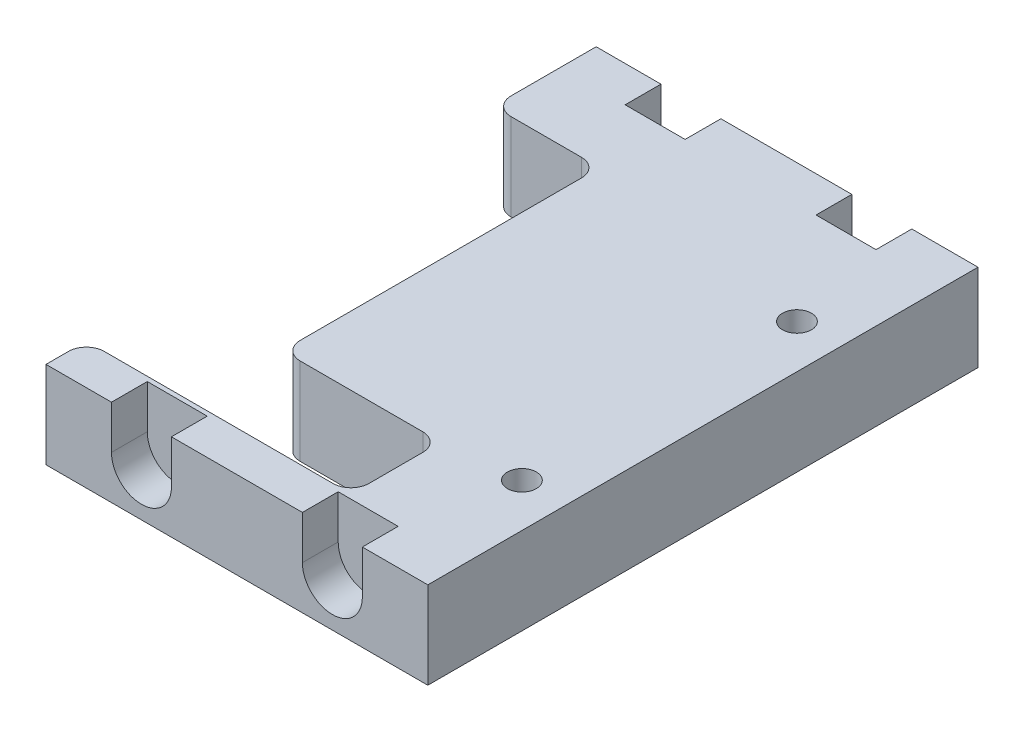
SolidWorks part; units mm, degrees
ref_plane "Front Plane" through (0, 0, 0) normal (0, 0, 1) x (1, 0, 0)
ref_plane "Top Plane" through (0, 0, 0) normal (0, 1, 0) x (1, 0, 0)
ref_plane "Right Plane" through (0, 0, 0) normal (1, 0, 0) x (0, 0, -1)
sketch "Sketch1" plane through (0, 0, 0) normal (0, 0, 1) x (1, 0, 0)
  line L6 (-810.8141, 612.9135) -> (-817.6657, 612.9135)
  line L7 (-810.8141, 612.9135) -> (-779.225, 612.9135)
  line L8 (-493.7649, 564.4955) -> (-493.7649, 1167.7963)
  line L9 (-493.7649, 1167.7963) -> (-817.6657, 1167.7963)
  line L10 (-817.6657, 1167.7963) -> (-817.6657, 564.4955)
  line L11 (-817.6657, 564.4955) -> (-493.7649, 564.4955)
  line L12 (-779.225, 612.9135) -> (-779.225, 571.3471)
  line L13 (-779.225, 571.3471) -> (-779.225, 564.4955)
  circle A2 centre (-798.6157, 583.5455) radius 2.667
extrude "Boss-Extrude1" add sketch "Sketch1" along normal blind 6.35 contours L13 L12 L7 L6 L10 L11 A2
sketch "Sketch2" plane through (0, 0, 6.35) normal (0, 0, 1) x (1, 0, 0)
  line L0 (-779.225, 564.4955) -> (-779.225, 555.0975)
  line L1 (-817.6657, 612.9135) -> (-827.0637, 612.9135)
  line L3 (-827.0637, 612.9135) -> (-779.225, 612.9135)
  line L4 (-779.225, 564.4955) -> (-779.225, 612.9135)
  line L5 (-779.225, 612.9135) -> (-817.6657, 612.9135)
  line L6 (-817.6657, 612.9135) -> (-817.6657, 564.4955)
  line L7 (-817.6657, 564.4955) -> (-779.225, 564.4955)
  line L8 (-779.225, 564.4955) -> (-779.225, 612.9135)
  line L9 (-779.225, 612.9135) -> (-817.6657, 612.9135)
  line L10 (-817.6657, 612.9135) -> (-817.6657, 564.4955)
  line L11 (-817.6657, 564.4955) -> (-779.225, 564.4955)
  line L12 (-827.0637, 612.9135) -> (-827.0637, 555.0975)
  line L13 (-827.0637, 555.0975) -> (-779.225, 555.0975)
  line L14 (-779.225, 612.9135) -> (-779.225, 555.0975)
  dimension "D2" = 9.398
  dimension "D1" = 0
extrude "Boss-Extrude2" add sketch "Sketch2" against normal up to vertex (996.0964 mm away) contours L12 L13 L0 L1 M15 M14
sketch "Sketch6" plane through (0, 0, 0) normal (0, 0, -1) x (-1, 0, 0)
  line L4 (779.225, 612.9135) -> (779.225, 555.0975)
  line L5 (779.225, 555.0975) -> (827.0637, 555.0975)
  line L6 (827.0637, 555.0975) -> (827.0637, 612.9135)
  line L7 (827.0637, 612.9135) -> (779.225, 612.9135)
  line L8 (779.225, 612.9135) -> (779.225, 555.0975)
  line L9 (779.225, 555.0975) -> (827.0637, 555.0975)
  line L10 (827.0637, 555.0975) -> (827.0637, 612.9135)
  line L11 (827.0637, 612.9135) -> (779.225, 612.9135)
  line L12 (804.9657, 562.1587) -> (817.4117, 562.1587)
  line L14 (819.1897, 562.1587) -> (820.0025, 562.1587)
  line L15 (820.0025, 562.1587) -> (820.0025, 612.9135)
  line L20 (817.4117, 562.1587) -> (819.1897, 562.1587)
  line L21 (804.9657, 562.1587) -> (779.225, 562.1587)
  dimension "D1" = 0
extrude "Boss-Extrude4" add sketch "Sketch6" along normal up to surface (78.0796 mm away) contours L12 L21 L8 L15 L14 L20 M11 M12 M13
sketch "Sketch7" plane through (0, 0, -78.0796) normal (0, 0, -1) x (-1, 0, 0)
  line L6 (805.2197, 576.9415) -> (805.2197, 612.9135)
  line L7 (779.225, 576.9415) -> (804.6609, 576.9415)
  line L8 (820.0025, 612.9135) -> (827.0637, 612.9135)
  line L9 (827.0637, 612.9135) -> (827.0637, 555.0975)
  line L10 (827.0637, 555.0975) -> (779.225, 555.0975)
  line L11 (779.225, 555.0975) -> (779.225, 562.1587)
  line L12 (779.225, 562.1587) -> (779.225, 576.9415)
  line L13 (820.0025, 612.9135) -> (805.2197, 612.9135)
  line L14 (804.6609, 576.9415) -> (805.2197, 576.9415)
  circle A2 centre (791.9609, 571.3471) radius 2.3812
  circle A3 centre (810.8141, 600.2587) radius 2.3812
sketch "Sketch8" plane through (0, 0, -78.0796) normal (0, 0, -1) x (-1, 0, 0)
  line L9 (805.2197, 612.9135) -> (805.2197, 576.9415)
  line L10 (820.0025, 612.9135) -> (805.2197, 612.9135)
  line L11 (827.0637, 612.9135) -> (820.0025, 612.9135)
  line L12 (827.0637, 555.0975) -> (827.0637, 612.9135)
  line L13 (779.225, 555.0975) -> (827.0637, 555.0975)
  line L14 (779.225, 562.1587) -> (779.225, 555.0975)
  line L15 (779.225, 576.9415) -> (779.225, 562.1587)
  line L16 (804.6609, 576.9415) -> (779.225, 576.9415)
  line L17 (805.2197, 576.9415) -> (804.6609, 576.9415)
  line L18 (805.2197, 612.9135) -> (805.2197, 576.9415)
  line L19 (820.0025, 612.9135) -> (805.2197, 612.9135)
  line L20 (827.0637, 612.9135) -> (820.0025, 612.9135)
  line L21 (827.0637, 555.0975) -> (827.0637, 612.9135)
  line L22 (779.225, 555.0975) -> (827.0637, 555.0975)
  line L23 (779.225, 562.1587) -> (779.225, 555.0975)
  line L24 (779.225, 576.9415) -> (779.225, 562.1587)
  line L25 (804.6609, 576.9415) -> (779.225, 576.9415)
  line L26 (805.2197, 576.9415) -> (804.6609, 576.9415)
  circle A1 centre (810.8141, 600.2587) radius 2.3813
  circle A2 centre (810.8141, 600.2587) radius 2.3812
  circle A3 centre (791.9609, 571.3471) radius 2.3813
  circle A4 centre (791.9609, 571.3471) radius 2.3812
  dimension "D1" = 0
  dimension "D2" = 0
  dimension "D3" = 0
extrude "Boss-Extrude6" add sketch "Sketch8" along normal blind 2.54
other "Cavity1"
other "5 SIDED ENCLOSURE 3 INCH.stp<1>@Assem11"
sketch "Sketch9" plane through (0, 612.9135, 0) normal (0, 1, 0) x (1, 0, 0)
  line L0 (-820.7645, 76.454) -> (-820.8153, 73.0504)
  line L1 (-820.8153, 3.1496) -> (-820.8153, 0)
  line L2 (-820.8153, 0) -> (-820.0025, 0)
  line L3 (-820.0025, 76.454) -> (-820.0025, 78.0796)
  line L4 (-820.0025, 78.0796) -> (-820.0025, 0)
  line L5 (-820.8153, 0) -> (-821.0693, 0)
  line L6 (-821.0693, 0) -> (-821.0693, 78.0796)
  line L7 (-821.0693, 78.0796) -> (-820.7645, 78.0796)
  line L12 (-820.7645, 76.454) -> (-820.7645, 78.0796)
  line L13 (-820.7645, 78.0796) -> (-805.2197, 78.0796)
  line L14 (-805.2197, 78.0796) -> (-805.2197, 80.6196)
  line L15 (-805.2197, 80.6196) -> (-827.0637, 80.6196)
  line L16 (-827.0637, 80.6196) -> (-827.0637, -6.35)
  line L17 (-827.0637, -6.35) -> (-779.225, -6.35)
  line L18 (-779.225, -6.35) -> (-779.225, 0)
  line L19 (-779.225, 0) -> (-820.0025, 0)
  line L20 (-820.0025, 0) -> (-820.0025, 1.0379)
  line L21 (-820.8153, 3.1496) -> (-820.8153, 73.0504)
  line L22 (-820.0025, 75.1621) -> (-820.0025, 76.454)
  line L23 (-820.0025, 76.454) -> (-820.7645, 76.454)
  line L24 (-820.7645, 76.454) -> (-820.7645, 78.0796)
  line L25 (-820.7645, 78.0796) -> (-805.2197, 78.0796)
  line L26 (-805.2197, 78.0796) -> (-805.2197, 80.6196)
  line L27 (-805.2197, 80.6196) -> (-827.0637, 80.6196)
  line L28 (-827.0637, 80.6196) -> (-827.0637, -6.35)
  line L29 (-827.0637, -6.35) -> (-779.225, -6.35)
  line L30 (-779.225, -6.35) -> (-779.225, 0)
  line L31 (-779.225, 0) -> (-820.0025, 0)
  line L32 (-820.0025, 0) -> (-820.0025, 1.0379)
  line L33 (-820.8153, 3.1496) -> (-820.8153, 73.0504)
  line L34 (-820.0025, 75.1621) -> (-820.0025, 76.454)
  line L35 (-820.0025, 76.454) -> (-820.7645, 76.454)
  arc A2 (-820.8153, 3.1496) -> (-820.0025, 1.0379) centre (-817.6657, 3.1496) ccw
  arc A3 (-820.0025, 75.1621) -> (-820.8153, 73.0504) centre (-817.6657, 73.0504) ccw
  arc A4 (-820.8153, 3.1496) -> (-820.0025, 1.0379) centre (-817.6657, 3.1496) ccw
  arc A5 (-820.0025, 75.1621) -> (-820.8153, 73.0504) centre (-817.6657, 73.0504) ccw
  dimension "D2" = 0.254
  dimension "D1" = 0
extrude "Cut-Extrude3" cut sketch "Sketch9" against normal up to surface (50.7548 mm away) contours L0 M28 M26 M27 | L7 L6 L5 L1 L0 M25 M26 M15 | L1 L2 M23 M24
sketch "Sketch10" plane through (-779.225, 0, 0) normal (1, 0, 0) x (0, 0, -1)
  line L0 (78.0796, 561.3459) -> (78.0796, 561.0919)
  line L1 (78.0796, 561.0919) -> (0, 561.0919)
  line L2 (0, 561.0919) -> (0, 562.1587)
  line L4 (24.4475, 562.1587) -> (24.4475, 561.3459) construction
  line L5 (24.4475, 562.1587) -> (24.4475, 561.3459)
  line L6 (0, 562.4127) -> (0, 562.1587)
  line L7 (0, 562.4127) -> (78.0796, 562.4127)
  line L8 (76.1963, 562.4127) -> (76.1963, 562.1587)
  line L9 (78.0796, 562.4127) -> (76.1963, 562.4127)
  line L10 (78.0796, 562.4127) -> (78.0796, 565.7277)
  line L11 (78.0796, 565.7277) -> (76.1963, 565.7277)
  line L12 (78.0796, 576.9415) -> (78.0796, 561.3459)
  line L13 (78.0796, 561.3459) -> (76.454, 561.3459)
  line L14 (76.454, 561.3459) -> (76.454, 562.1587)
  line L15 (76.454, 562.1587) -> (75.1621, 562.1587)
  line L16 (73.0504, 561.3459) -> (3.1496, 561.3459)
  line L17 (1.0379, 562.1587) -> (0, 562.1587)
  line L18 (0, 562.1587) -> (0, 612.9135)
  line L19 (0, 612.9135) -> (-6.35, 612.9135)
  line L20 (-6.35, 612.9135) -> (-6.35, 555.0975)
  line L21 (-6.35, 555.0975) -> (80.6196, 555.0975)
  line L22 (80.6196, 555.0975) -> (80.6196, 576.9415)
  line L23 (80.6196, 576.9415) -> (78.0796, 576.9415)
  line L24 (78.0796, 576.9415) -> (78.0796, 561.3459)
  line L25 (78.0796, 561.3459) -> (76.454, 561.3459)
  line L26 (76.454, 561.3459) -> (76.454, 562.1587)
  line L27 (76.454, 562.1587) -> (75.1621, 562.1587)
  line L28 (73.0504, 561.3459) -> (3.1496, 561.3459)
  line L29 (1.0379, 562.1587) -> (0, 562.1587)
  line L30 (0, 562.1587) -> (0, 612.9135)
  line L31 (0, 612.9135) -> (-6.35, 612.9135)
  line L32 (-6.35, 612.9135) -> (-6.35, 555.0975)
  line L33 (-6.35, 555.0975) -> (80.6196, 555.0975)
  line L34 (80.6196, 555.0975) -> (80.6196, 576.9415)
  line L35 (80.6196, 576.9415) -> (78.0796, 576.9415)
  line L36 (76.1963, 562.4127) -> (76.1963, 565.7277)
  line L37 (0, 561.0919) -> (3.4229, 561.0919)
  line L38 (0, 561.0919) -> (0, 564.0863)
  line L39 (0, 564.0863) -> (3.4229, 564.0863)
  line L40 (3.4229, 561.0919) -> (3.4229, 564.0863)
  arc A2 (73.0504, 561.3459) -> (75.1621, 562.1587) centre (73.0504, 564.4955) ccw
  arc A3 (1.0379, 562.1587) -> (3.1496, 561.3459) centre (3.1496, 564.4955) ccw
  arc A4 (73.0504, 561.3459) -> (75.1621, 562.1587) centre (73.0504, 564.4955) ccw
  arc A5 (1.0379, 562.1587) -> (3.1496, 561.3459) centre (3.1496, 564.4955) ccw
  dimension "D2" = 0.254
  dimension "D3" = 0.254
  dimension "D1" = 0
extrude "Cut-Extrude5" cut sketch "Sketch10" against normal up to surface (41.8444 mm away)
sketch "Sketch12" plane through (0, 0, -80.6196) normal (0, 0, -1) x (-1, 0, 0)
  line L6 (827.0637, 612.9135) -> (805.2197, 612.9135)
  line L7 (805.2197, 612.9135) -> (805.2197, 576.9415)
  line L8 (805.2197, 576.9415) -> (779.225, 576.9415)
  line L9 (779.225, 576.9415) -> (779.225, 555.0975)
  line L10 (779.225, 555.0975) -> (827.0637, 555.0975)
  line L11 (827.0637, 555.0975) -> (827.0637, 612.9135)
  line L12 (827.0637, 612.9135) -> (805.2197, 612.9135)
  line L13 (805.2197, 612.9135) -> (805.2197, 576.9415)
  line L14 (805.2197, 576.9415) -> (779.225, 576.9415)
  line L15 (779.225, 576.9415) -> (779.225, 555.0975)
  line L16 (779.225, 555.0975) -> (827.0637, 555.0975)
  line L17 (827.0637, 555.0975) -> (827.0637, 612.9135)
  circle A1 centre (791.9609, 571.3471) radius 2.3813
  circle A2 centre (791.9609, 571.3471) radius 2.3812
  circle A3 centre (810.8141, 600.2587) radius 2.3813
  circle A4 centre (810.8141, 600.2587) radius 2.3812
  dimension "D1" = 0
  dimension "D2" = 0
  dimension "D3" = 0
extrude "Boss-Extrude7" add sketch "Sketch12" along normal blind 3.81
sketch "Sketch13" plane through (0, 0, -84.4296) normal (0, 0, -1) x (-1, 0, 0)
  line L0 (797.5235, 571.3471) -> (797.5235, 576.9415)
  line L1 (805.2197, 576.9415) -> (779.225, 576.9415) construction
  line L2 (786.3983, 571.3471) -> (786.3983, 576.9415)
  line L3 (810.8141, 594.6961) -> (805.2197, 594.6961)
  line L4 (805.2197, 612.9135) -> (805.2197, 576.9415) construction
  line L5 (810.8141, 605.8213) -> (805.2197, 605.8213)
  line L12 (827.0637, 612.9135) -> (805.2197, 612.9135)
  line L13 (805.2197, 612.9135) -> (805.2197, 576.9415)
  line L14 (805.2197, 576.9415) -> (779.225, 576.9415)
  line L15 (779.225, 576.9415) -> (779.225, 555.0975)
  line L16 (779.225, 555.0975) -> (827.0637, 555.0975)
  line L17 (827.0637, 555.0975) -> (827.0637, 612.9135)
  line L18 (827.0637, 612.9135) -> (805.2197, 612.9135)
  line L19 (805.2197, 612.9135) -> (805.2197, 576.9415)
  line L20 (805.2197, 576.9415) -> (779.225, 576.9415)
  line L21 (779.225, 576.9415) -> (779.225, 555.0975)
  line L22 (779.225, 555.0975) -> (827.0637, 555.0975)
  line L23 (827.0637, 555.0975) -> (827.0637, 612.9135)
  circle A2 centre (810.8141, 600.2587) radius 3.0226
  circle A3 centre (791.9609, 571.3471) radius 3.0226
  circle A4 centre (791.9609, 571.3471) radius 5.5626
  circle A5 centre (810.8141, 600.2587) radius 5.5626
  dimension "D1" = 2.54
  dimension "D2" = 0
extrude "Cut-Extrude7" cut sketch "Sketch13" against normal blind 5.715 contours M16 | A5 A2 | A5 L5 L3 M7 | M3 | A3 M3 | A4 A3 | A4 L0 L2 M9
fillet "Fillet3" radius 1.27 4 edges at (-805.2197, 605.8213, -81.5721) (-805.2197, 594.6961, -81.5721) (-797.5235, 576.9415, -81.5721) (-786.3983, 576.9415, -81.5721)
sketch "Sketch14" plane through (0, 0, 6.35) normal (0, 0, 1) x (1, 0, 0)
  line L4 (-779.225, 612.9135) -> (-827.0637, 612.9135)
  line L5 (-827.0637, 612.9135) -> (-827.0637, 555.0975)
  line L6 (-827.0637, 555.0975) -> (-779.225, 555.0975)
  line L7 (-779.225, 555.0975) -> (-779.225, 612.9135)
  line L8 (-779.225, 612.9135) -> (-827.0637, 612.9135)
  line L9 (-827.0637, 612.9135) -> (-827.0637, 555.0975)
  line L10 (-827.0637, 555.0975) -> (-779.225, 555.0975)
  line L11 (-779.225, 555.0975) -> (-779.225, 612.9135)
  circle A1 centre (-798.6157, 583.5455) radius 12.7
  circle A2 centre (-798.6157, 583.5455) radius 12.954
  dimension "D1" = 0
  dimension "D2" = 0.254
extrude "Cut-Extrude8" cut sketch "Sketch14" against normal blind 5.715 contours A2 A1 | A1 M9 | M9
fillet "Fillet4" radius 2.54 3 edges at (-779.225, 576.9415, -81.2546) (-805.2197, 612.9135, -81.2546) (-779.225, 612.9135, 3.175)
sketch "Sketch15" plane through (0, 612.9135, 0) normal (0, 1, 0) x (1, 0, 0)
  line L4 (-827.0637, -6.35) -> (-779.225, -6.35)
  line L5 (-827.0637, 84.4296) -> (-827.0637, -6.35)
  line L6 (-779.225, 84.4296) -> (-827.0637, 84.4296)
  line L7 (-779.225, -6.35) -> (-779.225, 84.4296)
  line L8 (-827.0637, -6.35) -> (-779.225, -6.35)
  line L9 (-827.0637, 84.4296) -> (-827.0637, -6.35)
  line L10 (-779.225, 84.4296) -> (-827.0637, 84.4296)
  line L11 (-779.225, -6.35) -> (-779.225, 84.4296)
  dimension "D1" = 0
extrude "Cut-Extrude9" cut sketch "Sketch15" against normal up to surface (51.8216 mm away)
sketch "Sketch16" plane through (0, 555.0975, 0) normal (0, -1, 0) x (1, 0, 0)
  line L4 (-779.225, 6.35) -> (-827.0637, 6.35)
  line L5 (-827.0637, 6.35) -> (-827.0637, -84.4296)
  line L6 (-827.0637, -84.4296) -> (-779.225, -84.4296)
  line L7 (-779.225, -84.4296) -> (-779.225, 6.35)
  line L8 (-779.225, 6.35) -> (-827.0637, 6.35)
  line L9 (-827.0637, 6.35) -> (-827.0637, -84.4296)
  line L10 (-827.0637, -84.4296) -> (-779.225, -84.4296)
  line L11 (-779.225, -84.4296) -> (-779.225, 6.35)
  dimension "D1" = 0
extrude "Boss-Extrude8" add sketch "Sketch16" along normal blind 6.35
sketch "Sketch17" plane through (-827.0637, 0, 0) normal (-1, 0, 0) x (0, 0, 1)
  line L4 (6.35, 548.7475) -> (6.35, 561.0919)
  line L5 (6.35, 561.0919) -> (-84.4296, 561.0919)
  line L6 (-84.4296, 561.0919) -> (-84.4296, 548.7475)
  line L7 (-84.4296, 548.7475) -> (6.35, 548.7475)
  line L8 (6.35, 548.7475) -> (6.35, 561.0919)
  line L9 (6.35, 561.0919) -> (-84.4296, 561.0919)
  line L10 (-84.4296, 561.0919) -> (-84.4296, 548.7475)
  line L11 (-84.4296, 548.7475) -> (6.35, 548.7475)
  dimension "D1" = 0
extrude "Boss-Extrude9" add sketch "Sketch17" along normal up to surface (6.35 mm away)
other "Cavity2"
other "Bottom<1>@Bumper Assembly1"
other "Top<1>@Bumper Assembly1"
other "Cavity3"
other "Long Side<1>@Bumper Assembly1"
sketch "Sketch18" plane through (0, 548.7475, 0) normal (0, -1, 0) x (1, 0, 0)
  line L0 (-782.4, -48.26) -> (-830.2387, -48.26) construction
  line L5 (-806.3194, -84.4296) -> (-806.3194, -10.16) construction
  line L6 (-782.4, -60.96) -> (-830.2387, -60.96) construction
  line L7 (-833.4137, -84.4296) -> (-779.225, -84.4296) construction
  line L14 (-833.4137, -84.4296) -> (-779.225, -84.4296) construction
  line L21 (-779.225, -84.4296) -> (-833.4137, 6.35) construction
  line L22 (-779.225, 6.35) -> (-833.4137, 6.35) construction
  line L27 (-782.4, -35.56) -> (-830.2387, -35.56) construction
  line L28 (-782.4, -22.86) -> (-830.2387, -22.86) construction
  line L29 (-782.4, -10.16) -> (-830.2387, -10.16) construction
  text T0 "<b>R</b>" font "Century Gothic" height in points 36
  text T1 "I" font "Century Gothic" height in points 36
  text T2 "F" font "Century Gothic" height in points 36
  text T3 "T" font "Century Gothic" height in points 36
  text T4 "S" font "Century Gothic" height in points 36
  point P1 (-806.3194, -84.4296)
  point P15 (-806.3194, -60.96)
  point P27 (-806.3194, -39.0398)
  dimension "D2" = 16.51
  dimension "D1" = 12.7
  dimension "D4" = 5
extrude "Cut-Extrude10" cut sketch "Sketch18" against normal through all
sketch "Sketch19" plane through (0, 548.7475, 0) normal (0, -1, 0) x (1, 0, 0)
  line L3 (-805.8633, -68.7754) -> (-805.2814, -68.7754)
  line L4 (-805.2814, -68.7754) -> (-805.2814, -66.8215)
  line L5 (-805.2814, -66.8215) -> (-805.9473, -66.8215)
  line L6 (-805.8633, -68.7754) -> (-805.2814, -68.7754)
  line L7 (-805.2814, -68.7754) -> (-805.2814, -66.8215)
  line L8 (-805.2814, -66.8215) -> (-805.9473, -66.8215)
  spline S2 degree 3 poles (-791.841, 1933.0183) (-785.8141, -82.8061) (-796.1442, -66.4595) (-806.4088, -66.8324) (-806.6124, -66.852) (-806.7963, -66.8768) (-806.9615, -66.9054) (-807.1064, -66.9464) (-807.2333, -66.9903) (-807.3405, -67.0451) (-807.4325, -67.1064) (-807.5095, -67.179) (-807.5774, -67.2586) (-807.6307, -67.3501) (-807.6737, -67.4498) (-807.7004, -67.5596) (-808.3447, -71.1457) (-783.6708, -77.0657) (-2799.9016, 108.2283) knots -13.020716 -13.020716 -13.020716 -13.020716 0.105558 0.202122 0.290736 0.370617 0.442748 0.507764 0.565672 0.616562 0.663447 0.708377 0.753458 0.798569 0.845127 0.893728 0.944698 5.557546 5.557546 5.557546 5.557546 only from (-805.9473, -66.8215) to (-807.7237, -67.8023)
  spline S3 degree 3 poles (-2791.4355, -321.8292) (-779.4289, -57.0269) (-808.6486, -64.5495) (-807.6793, -68.0937) (-807.6206, -68.2264) (-807.5374, -68.3477) (-807.4337, -68.4537) (-807.3148, -68.5467) (-807.1785, -68.6211) (-807.0526, -68.6718) (-806.9363, -68.701) (-806.8319, -68.722) (-806.7109, -68.7389) (-806.5733, -68.7514) (-806.4194, -68.7632) (-806.2488, -68.7706) (-793.917, -68.9867) (-781.5432, -57.7566) (-786.6414, -2068.5426) knots -4.428971 -4.428971 -4.428971 -4.428971 0.063753 0.124452 0.185322 0.2467 0.3093 0.372394 0.436875 0.505164 0.543418 0.588552 0.639762 0.697972 0.76333 0.83502 0.913895 16.367288 16.367288 16.367288 16.367288 only from (-807.7237, -67.8023) to (-805.8633, -68.7754)
  spline S4 degree 3 poles (-805.9473, -66.8215) (-806.0287, -66.8225) (-806.1846, -66.8242) (-806.4088, -66.8324) (-806.6124, -66.852) (-806.7963, -66.8768) (-806.9615, -66.9054) (-807.1064, -66.9464) (-807.2333, -66.9903) (-807.3405, -67.0451) (-807.4325, -67.1064) (-807.5095, -67.179) (-807.5774, -67.2586) (-807.6307, -67.3501) (-807.6737, -67.4498) (-807.7004, -67.5596) (-807.7216, -67.6775) (-807.723, -67.7596) (-807.7237, -67.8023) knots 0 0 0 0 0.105558 0.202122 0.290736 0.370617 0.442748 0.507764 0.565672 0.616562 0.663447 0.708377 0.753458 0.798569 0.845127 0.893728 0.944698 1 1 1 1
  spline S5 degree 3 poles (-807.7237, -67.8023) (-807.7219, -67.8528) (-807.7183, -67.9514) (-807.6793, -68.0937) (-807.6206, -68.2264) (-807.5374, -68.3477) (-807.4337, -68.4537) (-807.3148, -68.5467) (-807.1785, -68.6211) (-807.0526, -68.6718) (-806.9363, -68.701) (-806.8319, -68.722) (-806.7109, -68.7389) (-806.5733, -68.7514) (-806.4194, -68.7632) (-806.2488, -68.7706) (-806.0618, -68.7739) (-805.9314, -68.7749) (-805.8633, -68.7754) knots 0 0 0 0 0.063753 0.124452 0.185322 0.2467 0.3093 0.372394 0.436875 0.505164 0.543418 0.588552 0.639762 0.697972 0.76333 0.83502 0.913895 1 1 1 1
  dimension "D1" = 0
extrude "Cut-Extrude11" cut sketch "Sketch19" against normal up to surface (12.3444 mm away)
ref_plane "Plane1" through (-776.685, 0, 0) normal (1, 0, 0) x (0, 0, -1)
mirror "Mirror1" about plane through (-776.685, 0, 0) normal (1, 0, 0)
sketch "Sketch20" plane through (0, 548.7475, 0) normal (0, -1, 0) x (1, 0, 0)
  line L4 (-779.225, -84.4296) -> (-779.225, 6.35)
  line L5 (-779.225, 6.35) -> (-833.4137, 6.35)
  line L6 (-833.4137, 6.35) -> (-833.4137, -84.4296)
  line L7 (-833.4137, -84.4296) -> (-779.225, -84.4296)
  line L8 (-779.225, -84.4296) -> (-779.225, 6.35)
  line L9 (-779.225, 6.35) -> (-833.4137, 6.35)
  line L10 (-833.4137, 6.35) -> (-833.4137, -84.4296)
  line L11 (-833.4137, -84.4296) -> (-779.225, -84.4296)
  dimension "D1" = 0
extrude "Cut-Extrude12" cut sketch "Sketch20" against normal through all
sketch "Sketch21" plane through (0, 554.8689, 0) normal (0, 1, 0) x (1, 0, 0)
  line L4 (-726.3062, 84.4296) -> (-726.3062, -6.35)
  line L5 (-726.3062, -6.35) -> (-719.9562, -6.35)
  line L6 (-719.9562, -6.35) -> (-719.9562, 84.4296)
  line L7 (-719.9562, 84.4296) -> (-726.3062, 84.4296)
  line L8 (-726.3062, 84.4296) -> (-726.3062, -6.35)
  line L9 (-726.3062, -6.35) -> (-719.9562, -6.35)
  line L10 (-719.9562, -6.35) -> (-719.9562, 84.4296)
  line L11 (-719.9562, 84.4296) -> (-726.3062, 84.4296)
  dimension "D1" = 0
extrude "Boss-Extrude10" add sketch "Sketch21" along normal up to surface (0.2286 mm away)
sketch "Sketch22" plane through (0, 548.7475, 0) normal (0, -1, 0) x (1, 0, 0)
  line L2 (-750.1035, -11.944) -> (-748.5999, -12.8465)
  line L3 (-744.4862, -18.4123) -> (-745.7646, -17.2427)
  line L4 (-746.3179, -48.26) -> (-748.0275, -48.26)
  line L5 (-746.3179, -57.785) -> (-746.3179, -48.26)
  line L6 (-748.0275, -57.785) -> (-746.3179, -57.785)
  line L7 (-748.0275, -48.26) -> (-748.0275, -57.785)
  line L8 (-748.0886, -60.96) -> (-749.7982, -60.96)
  line L9 (-748.0886, -65.1119) -> (-748.0886, -60.96)
  line L10 (-747.5085, -65.1119) -> (-748.0886, -65.1119)
  line L11 (-745.4097, -60.96) -> (-747.5085, -65.1119)
  line L12 (-743.5093, -60.96) -> (-745.4097, -60.96)
  line L13 (-745.7073, -65.3065) -> (-743.5093, -60.96)
  line L14 (-749.7982, -70.485) -> (-747.8062, -70.485)
  line L15 (-749.7982, -60.96) -> (-749.7982, -70.485)
  line L16 (-748.0886, -60.96) -> (-749.7982, -60.96)
  line L17 (-748.0886, -65.1119) -> (-748.0886, -60.96)
  line L18 (-747.5085, -65.1119) -> (-748.0886, -65.1119)
  line L19 (-745.4097, -60.96) -> (-747.5085, -65.1119)
  line L20 (-743.5093, -60.96) -> (-745.4097, -60.96)
  line L21 (-745.7073, -65.3065) -> (-743.5093, -60.96)
  line L22 (-749.7982, -70.485) -> (-747.8062, -70.485)
  line L23 (-749.7982, -60.96) -> (-749.7982, -70.485)
  line L24 (-746.3179, -48.26) -> (-748.0275, -48.26)
  line L25 (-746.3179, -57.785) -> (-746.3179, -48.26)
  line L26 (-748.0275, -57.785) -> (-746.3179, -57.785)
  line L27 (-748.0275, -48.26) -> (-748.0275, -57.785)
  line L28 (-750.1035, -11.944) -> (-748.5999, -12.8465)
  line L29 (-744.4862, -18.4123) -> (-745.7646, -17.2427)
  line L32 (-747.9665, -30.6754) -> (-749.6761, -30.6754)
  line L33 (-747.9665, -22.86) -> (-747.9665, -30.6754)
  line L34 (-747.417, -35.56) -> (-749.1266, -35.56)
  line L35 (-747.417, -39.834) -> (-747.417, -35.56)
  line L36 (-744.4862, -39.834) -> (-747.417, -39.834)
  line L37 (-744.4862, -41.5437) -> (-744.4862, -39.834)
  line L38 (-747.417, -41.5437) -> (-744.4862, -41.5437)
  line L39 (-747.417, -43.3754) -> (-747.417, -41.5437)
  line L40 (-744.4862, -43.3754) -> (-747.417, -43.3754)
  line L41 (-744.4862, -45.085) -> (-744.4862, -43.3754)
  line L42 (-749.1266, -45.085) -> (-744.4862, -45.085)
  line L43 (-749.1266, -35.56) -> (-749.1266, -45.085)
  line L44 (-747.417, -35.56) -> (-749.1266, -35.56)
  line L45 (-747.417, -39.834) -> (-747.417, -35.56)
  line L46 (-744.4862, -39.834) -> (-747.417, -39.834)
  line L47 (-744.4862, -41.5437) -> (-744.4862, -39.834)
  line L48 (-747.417, -41.5437) -> (-744.4862, -41.5437)
  line L49 (-747.417, -43.3754) -> (-747.417, -41.5437)
  line L50 (-744.4862, -43.3754) -> (-747.417, -43.3754)
  line L51 (-744.4862, -45.085) -> (-744.4862, -43.3754)
  line L52 (-749.1266, -45.085) -> (-744.4862, -45.085)
  line L53 (-749.1266, -35.56) -> (-749.1266, -45.085)
  line L54 (-746.2569, -22.86) -> (-747.9665, -22.86)
  line L55 (-746.2569, -30.6754) -> (-746.2569, -22.86)
  line L56 (-744.5472, -30.6754) -> (-746.2569, -30.6754)
  line L57 (-744.5472, -32.385) -> (-744.5472, -30.6754)
  line L58 (-749.6761, -32.385) -> (-744.5472, -32.385)
  line L59 (-749.6761, -30.6754) -> (-749.6761, -32.385)
  line L60 (-747.9665, -30.6754) -> (-749.6761, -30.6754)
  line L61 (-747.9665, -22.86) -> (-747.9665, -30.6754)
  line L62 (-746.2569, -22.86) -> (-747.9665, -22.86)
  line L63 (-746.2569, -30.6754) -> (-746.2569, -22.86)
  line L64 (-744.5472, -30.6754) -> (-746.2569, -30.6754)
  line L65 (-744.5472, -32.385) -> (-744.5472, -30.6754)
  line L66 (-749.6761, -32.385) -> (-744.5472, -32.385)
  line L67 (-749.6761, -30.6754) -> (-749.6761, -32.385)
  spline S2 degree 3 poles (3253.275, 74.1316) (-777.0296, -87.0287) (-743.1812, -76.4884) (-743.9603, -67.3408) (-743.9945, -67.1334) (-744.0447, -66.9361) (-744.1048, -66.747) (-744.1826, -66.5691) (-744.2711, -66.3991) (-744.376, -66.2399) (-744.4912, -66.088) (-744.6251, -65.949) (-744.77, -65.8163) (-744.9303, -65.6944) (-745.1056, -65.584) (-745.2925, -65.4807) (-753.0233, -61.8543) (-775.2465, -93.9017) (743.44, 3646.85) knots -8.197893 -8.197893 -8.197893 -8.197893 0.068738 0.134783 0.198527 0.260938 0.320957 0.379897 0.438493 0.496142 0.55425 0.612731 0.672493 0.733974 0.796799 0.861942 0.929401 8.604127 8.604127 8.604127 8.604127 only from (-743.9367, -67.7794) to (-745.7073, -65.3065)
  spline S3 degree 3 poles (-712.7597, -4070.0176) (-779.4214, -36.678) (-762.9373, -71.0909) (-747.0561, -70.4694) (-746.7206, -70.45) (-746.414, -70.4186) (-746.1367, -70.3826) (-745.8891, -70.3342) (-745.6705, -70.2805) (-745.478, -70.2144) (-745.3048, -70.1385) (-745.1439, -70.0525) (-744.9914, -69.9541) (-744.8484, -69.8437) (-744.7105, -69.7255) (-744.585, -69.5925) (-744.4664, -69.4491) (-744.356, -69.2953) (-744.2568, -69.1315) (-744.1712, -68.9596) (-744.0976, -68.7807) (-744.0393, -68.5941) (-743.9928, -68.4003) (-743.9617, -68.1999) (-743.1235, -60.6665) (-782.8085, -50.9653) (3250.9611, -266.0624) knots -8.591711 -8.591711 -8.591711 -8.591711 0.072858 0.140126 0.202191 0.258785 0.31065 0.356897 0.398298 0.435139 0.469338 0.502878 0.535973 0.569621 0.602796 0.636402 0.67065 0.705713 0.741084 0.776499 0.811858 0.848034 0.884571 0.922007 0.960215 5.074251 5.074251 5.074251 5.074251 only from (-747.8062, -70.485) to (-743.9367, -67.7794)
  spline S4 degree 3 poles (-743.9367, -67.7794) (-743.9384, -67.7043) (-743.9419, -67.5571) (-743.9603, -67.3408) (-743.9945, -67.1334) (-744.0447, -66.9361) (-744.1048, -66.747) (-744.1826, -66.5691) (-744.2711, -66.3991) (-744.376, -66.2399) (-744.4912, -66.088) (-744.6251, -65.949) (-744.77, -65.8163) (-744.9303, -65.6944) (-745.1056, -65.584) (-745.2925, -65.4807) (-745.4937, -65.3863) (-745.6351, -65.3335) (-745.7073, -65.3065) knots 0 0 0 0 0.068738 0.134783 0.198527 0.260938 0.320957 0.379897 0.438493 0.496142 0.55425 0.612731 0.672493 0.733974 0.796799 0.861942 0.929401 1 1 1 1
  spline S5 degree 3 poles (-747.8062, -70.485) (-747.6745, -70.4845) (-747.4213, -70.4837) (-747.0561, -70.4694) (-746.7206, -70.45) (-746.414, -70.4186) (-746.1367, -70.3826) (-745.8891, -70.3342) (-745.6705, -70.2805) (-745.478, -70.2144) (-745.3048, -70.1385) (-745.1439, -70.0525) (-744.9914, -69.9541) (-744.8484, -69.8437) (-744.7105, -69.7255) (-744.585, -69.5925) (-744.4664, -69.4491) (-744.356, -69.2953) (-744.2568, -69.1315) (-744.1712, -68.9596) (-744.0976, -68.7807) (-744.0393, -68.5941) (-743.9928, -68.4003) (-743.9617, -68.1999) (-743.9386, -67.9923) (-743.9373, -67.8513) (-743.9367, -67.7794) knots 0 0 0 0 0.072858 0.140126 0.202191 0.258785 0.31065 0.356897 0.398298 0.435139 0.469338 0.502878 0.535973 0.569621 0.602796 0.636402 0.67065 0.705713 0.741084 0.776499 0.811858 0.848034 0.884571 0.922007 0.960215 1 1 1 1
  spline S18 degree 3 poles (-4738.905, -305.9343) (-706.306, 0.6997) (-750.7404, -10.3835) (-749.5726, -17.9921) (-749.5182, -18.2199) (-749.4399, -18.4393) (-749.335, -18.6478) (-749.211, -18.8487) (-749.0645, -19.0415) (-748.8966, -19.2218) (-748.7123, -19.3875) (-748.5157, -19.533) (-748.3087, -19.6559) (-748.0906, -19.7561) (-747.8617, -19.8343) (-747.622, -19.8895) (-739.1771, -21.0028) (-727.9792, 21.5395) (-981.6023, -4012.8319) knots -5.768343 -5.768343 -5.768343 -5.768343 0.063175 0.124462 0.184848 0.244577 0.304549 0.365432 0.427356 0.491896 0.556136 0.619244 0.681136 0.742463 0.804983 0.868247 0.932885 7.394715 7.394715 7.394715 7.394715 only from (-749.615, -17.5136) to (-747.1155, -19.9292)
  spline S19 degree 3 poles (-3309.5986, 3056.6722) (-695.6814, -10.6656) (-732.023, -0.7272) (-747.8975, -14.7609) (-748.1936, -15.0329) (-748.4551, -15.2881) (-748.6825, -15.5251) (-748.8786, -15.7418) (-749.0401, -15.9424) (-749.2075, -16.1819) (-749.3711, -16.4697) (-749.5101, -16.8176) (-751.6123, -24.9465) (-693.2528, -40.8236) (-4718.7128, 475.1467) knots -14.65106 -14.65106 -14.65106 -14.65106 0.11214 0.215231 0.309946 0.396015 0.473203 0.541905 0.602297 0.654875 0.748186 0.835255 0.918914 6.639965 6.639965 6.639965 6.639965 only from (-747.2147, -14.1707) to (-749.615, -17.5136)
  spline S20 degree 3 poles (3213.4385, -579.0677) (-790.4419, 3.5799) (-744.6437, -8.0689) (-746.0079, -12.8569) (-746.0817, -13.0203) (-746.1663, -13.1558) (-746.2546, -13.2687) (-746.3411, -13.3651) (-746.4436, -13.4738) (-746.5648, -13.5919) (-746.7022, -13.7216) (-746.8564, -13.8626) (-757.7725, -23.429) (-784.1581, -14.7776) (1817.798, -3083.0362) knots -6.709352 -6.709352 -6.709352 -6.709352 0.076338 0.155074 0.238325 0.327891 0.378865 0.43968 0.509886 0.588921 0.677472 0.775572 0.882649 21.081322 21.081322 21.081322 21.081322 only from (-745.9516, -12.5279) to (-747.2147, -14.1707)
  spline S21 degree 3 poles (-239.3817, 3955.8621) (-765.2815, -61.8263) (-752.4602, -10.1462) (-746.6155, -11.6884) (-746.4261, -11.7717) (-746.2633, -11.8928) (-746.125, -12.0309) (-746.0259, -12.1867) (-744.3487, -16.5306) (-797.2647, -31.1444) (3186.4157, 718.1825) knots -11.112171 -11.112171 -11.112171 -11.112171 0.141922 0.275349 0.405274 0.536299 0.66224 0.777967 0.88833 9.47252 9.47252 9.47252 9.47252 only from (-747.0392, -11.6254) to (-745.9516, -12.5279)
  spline S22 degree 3 poles (-4143.3921, 2102.1735) (-719.1934, -54.1648) (-754.1139, -20.3878) (-748.2577, -12.3165) (-748.0729, -12.1036) (-747.8795, -11.9303) (-747.6797, -11.794) (-747.4726, -11.6967) (-741.685, -10.0706) (-728.6327, -61.276) (-1280.4084, 3952.293) knots -13.915115 -13.915115 -13.915115 -13.915115 0.160458 0.307612 0.442139 0.566229 0.681222 0.789558 0.895029 9.282627 9.282627 9.282627 9.282627 only from (-748.5999, -12.8465) to (-747.0392, -11.6254)
  spline S23 degree 3 poles (-918.3362, 3986.0187) (-727.9692, -47.1014) (-738.6977, -9.0694) (-747.5827, -9.9435) (-747.8124, -9.9811) (-748.0334, -10.0355) (-748.2473, -10.1027) (-748.4517, -10.1903) (-748.6492, -10.2892) (-748.8393, -10.4039) (-749.0204, -10.5371) (-749.1977, -10.6836) (-749.3648, -10.8513) (-749.5283, -11.0342) (-749.6812, -11.2376) (-749.8316, -11.4553) (-755.5959, -21.1828) (-729.6165, -47.8871) (-4288.0136, 1853.7281) knots -6.774381 -6.774381 -6.774381 -6.774381 0.063568 0.125901 0.186289 0.24504 0.303437 0.361056 0.418329 0.475792 0.534074 0.593626 0.655051 0.718698 0.784919 0.853484 0.925163 9.602134 9.602134 9.602134 9.602134 only from (-747.1021, -9.9158) to (-750.1035, -11.944)
  spline S24 degree 3 poles (3245.8952, 262.8839) (-790.4838, -32.5287) (-743.0359, -20.51) (-744.288, -12.066) (-744.3465, -11.8017) (-744.4366, -11.5519) (-744.5473, -11.3138) (-744.6823, -11.0872) (-744.8474, -10.8774) (-745.0307, -10.6787) (-745.2366, -10.5004) (-745.4581, -10.3432) (-745.6954, -10.2105) (-745.9469, -10.1011) (-746.2157, -10.02) (-746.4975, -9.9586) (-756.0419, -8.7722) (-768.1402, -54.1255) (-547.55, 3984.8518) knots -5.589368 -5.589368 -5.589368 -5.589368 0.06519 0.127905 0.189015 0.248502 0.307556 0.366963 0.426931 0.48828 0.550044 0.611324 0.672163 0.734187 0.796953 0.862273 0.929637 7.307067 7.307067 7.307067 7.307067 only from (-744.242, -12.6271) to (-747.1021, -9.9158)
  spline S25 degree 3 poles (2264.9475, -2648.6747) (-794.2561, -1.4389) (-751.7021, -23.2532) (-744.7709, -14.2742) (-744.5964, -14.011) (-744.4612, -13.7488) (-744.3632, -13.4823) (-744.2919, -13.2077) (-742.9866, -4.4583) (-789.9889, 7.5667) (3247.4785, -265.4161) knots -13.376111 -13.376111 -13.376111 -13.376111 0.150802 0.289894 0.417473 0.534875 0.648075 0.762455 0.879852 11.388611 11.388611 11.388611 11.388611 only from (-745.2265, -14.8118) to (-744.242, -12.6271)
  spline S26 degree 3 poles (1815.4632, -3081.8353) (-858.2339, -104.7491) (-800.1155, -62.3511) (-746.005, -15.523) (-745.8139, -15.3554) (-745.6494, -15.2062) (-745.5067, -15.0813) (-745.392, -14.9732) (-740.4633, -10.303) (-749.0882, 8.1302) (2067.3529, -2857.7244) knots -129.787107 -129.787107 -129.787107 -129.787107 0.192953 0.366186 0.520459 0.655785 0.770623 0.865677 0.942674 13.133776 13.133776 13.133776 13.133776 only from (-746.4534, -15.9109) to (-745.2265, -14.8118)
  spline S27 degree 3 poles (-3825.0552, 2537.3882) (-735.0048, -42.1498) (-751.4053, -21.1194) (-747.58, -16.9455) (-747.4569, -16.8249) (-747.3101, -16.6804) (-747.1339, -16.5176) (-746.9324, -16.3317) (-724.4033, 3.3832) (-712.4436, 34.4968) (2020.1812, -2903.5452) knots -9.267262 -9.267262 -9.267262 -9.267262 0.059231 0.13713 0.233823 0.348656 0.483195 0.636695 0.809253 50.765023 50.765023 50.765023 50.765023 only from (-747.747, -17.1397) to (-746.4534, -15.9109)
  spline S28 degree 3 poles (-4709.5024, 533.4999) (-706.9184, -31.0254) (-748.9292, -21.1547) (-747.8676, -17.3592) (-746.1299, -13.3317) (-707.7748, -29.9652) (-4226.9894, 1956.2202) knots -23.194495 -23.194495 -23.194495 -23.194495 0.241881 0.487115 0.737838 26.946146 26.946146 26.946146 26.946146 only from (-747.9054, -17.5957) to (-747.747, -17.1397)
  spline S29 degree 3 poles (-1192.0902, -3993.2501) (-732.4343, 26.8215) (-742.6525, -19.3756) (-747.4424, -18.177) (-747.5761, -18.1168) (-747.6911, -18.0338) (-747.7836, -17.9345) (-747.8556, -17.8289) (-749.1172, -14.3539) (-704.6301, -3.1897) (-4693.5344, -673.7153) knots -12.969028 -12.969028 -12.969028 -12.969028 0.14802 0.285787 0.415605 0.546256 0.67037 0.784556 0.893342 10.616813 10.616813 10.616813 10.616813 only from (-747.1346, -18.2196) to (-747.9054, -17.5957)
  spline S30 degree 3 poles (2441.0194, -2434.364) (-768.6332, 22.9946) (-740.0341, -10.6161) (-746.095, -17.6667) (-746.2645, -17.837) (-746.4365, -17.9745) (-746.608, -18.0851) (-746.7826, -18.1615) (-751.7912, -19.5605) (-763.6876, 27.4456) (-193.3323, -3979.4665) knots -15.488966 -15.488966 -15.488966 -15.488966 0.162432 0.311848 0.448466 0.574275 0.689054 0.797558 0.900286 9.552408 9.552408 9.552408 9.552408 only from (-745.7646, -17.2427) to (-747.1346, -18.2196)
  spline S31 degree 3 poles (-384.0341, -4003.2014) (-769.3777, 30.9914) (-755.3186, -21.5644) (-746.4491, -19.8531) (-746.126, -19.7517) (-745.8648, -19.6323) (-745.6588, -19.513) (-745.5005, -19.4053) (-745.3382, -19.2817) (-745.1748, -19.1385) (-745.0042, -18.984) (-744.835, -18.8076) (-737.3371, -10.753) (-756.1613, 20.4675) (2273.0718, -2643.5339) knots -8.258385 -8.258385 -8.258385 -8.258385 0.106908 0.212971 0.319769 0.429097 0.485871 0.546571 0.611442 0.680224 0.75359 0.830757 0.913135 11.240903 11.240903 11.240903 11.240903 only from (-747.1155, -19.9292) to (-744.4862, -18.4123)
  spline S32 degree 3 poles (-749.615, -17.5136) (-749.613, -17.5952) (-749.6089, -17.7558) (-749.5726, -17.9921) (-749.5182, -18.2199) (-749.4399, -18.4393) (-749.335, -18.6478) (-749.211, -18.8487) (-749.0645, -19.0415) (-748.8966, -19.2218) (-748.7123, -19.3875) (-748.5157, -19.533) (-748.3087, -19.6559) (-748.0906, -19.7561) (-747.8617, -19.8343) (-747.622, -19.8895) (-747.3721, -19.9225) (-747.2021, -19.927) (-747.1155, -19.9292) knots 0 0 0 0 0.063175 0.124462 0.184848 0.244577 0.304549 0.365432 0.427356 0.491896 0.556136 0.619244 0.681136 0.742463 0.804983 0.868247 0.932885 1 1 1 1
  spline S33 degree 3 poles (-747.2147, -14.1707) (-747.3359, -14.2733) (-747.5686, -14.4702) (-747.8975, -14.7609) (-748.1936, -15.0329) (-748.4551, -15.2881) (-748.6825, -15.5251) (-748.8786, -15.7418) (-749.0401, -15.9424) (-749.2075, -16.1819) (-749.3711, -16.4697) (-749.5101, -16.8176) (-749.6, -17.165) (-749.6101, -17.3986) (-749.615, -17.5136) knots 0 0 0 0 0.11214 0.215231 0.309946 0.396015 0.473203 0.541905 0.602297 0.654875 0.748186 0.835255 0.918914 1 1 1 1
  spline S34 degree 3 poles (-745.9516, -12.5279) (-745.9547, -12.5822) (-745.9611, -12.6926) (-746.0079, -12.8569) (-746.0817, -13.0203) (-746.1663, -13.1558) (-746.2546, -13.2687) (-746.3411, -13.3651) (-746.4436, -13.4738) (-746.5648, -13.5919) (-746.7022, -13.7216) (-746.8564, -13.8626) (-747.029, -14.0139) (-747.1509, -14.1169) (-747.2147, -14.1707) knots 0 0 0 0 0.076338 0.155074 0.238325 0.327891 0.378865 0.43968 0.509886 0.588921 0.677472 0.775572 0.882649 1 1 1 1
  spline S35 degree 3 poles (-747.0392, -11.6254) (-746.965, -11.6284) (-746.8212, -11.6341) (-746.6155, -11.6884) (-746.4261, -11.7717) (-746.2633, -11.8928) (-746.125, -12.0309) (-746.0259, -12.1867) (-745.9616, -12.3532) (-745.9549, -12.4694) (-745.9516, -12.5279) knots 0 0 0 0 0.141922 0.275349 0.405274 0.536299 0.66224 0.777967 0.88833 1 1 1 1
  spline S36 degree 3 poles (-748.5999, -12.8465) (-748.5444, -12.75) (-748.438, -12.5651) (-748.2577, -12.3165) (-748.0729, -12.1036) (-747.8795, -11.9303) (-747.6797, -11.794) (-747.4726, -11.6967) (-747.2581, -11.6364) (-747.112, -11.6291) (-747.0392, -11.6254) knots 0 0 0 0 0.160458 0.307612 0.442139 0.566229 0.681222 0.789558 0.895029 1 1 1 1
  spline S37 degree 3 poles (-747.1021, -9.9158) (-747.1836, -9.9172) (-747.3449, -9.9201) (-747.5827, -9.9435) (-747.8124, -9.9811) (-748.0334, -10.0355) (-748.2473, -10.1027) (-748.4517, -10.1903) (-748.6492, -10.2892) (-748.8393, -10.4039) (-749.0204, -10.5371) (-749.1977, -10.6836) (-749.3648, -10.8513) (-749.5283, -11.0342) (-749.6812, -11.2376) (-749.8316, -11.4553) (-749.9722, -11.6926) (-750.0591, -11.859) (-750.1035, -11.944) knots 0 0 0 0 0.063568 0.125901 0.186289 0.24504 0.303437 0.361056 0.418329 0.475792 0.534074 0.593626 0.655051 0.718698 0.784919 0.853484 0.925163 1 1 1 1
  spline S38 degree 3 poles (-744.242, -12.6271) (-744.2437, -12.5309) (-744.247, -12.3422) (-744.288, -12.066) (-744.3465, -11.8017) (-744.4366, -11.5519) (-744.5473, -11.3138) (-744.6823, -11.0872) (-744.8474, -10.8774) (-745.0307, -10.6787) (-745.2366, -10.5004) (-745.4581, -10.3432) (-745.6954, -10.2105) (-745.9469, -10.1011) (-746.2157, -10.02) (-746.4975, -9.9586) (-746.7952, -9.9216) (-746.9984, -9.9177) (-747.1021, -9.9158) knots 0 0 0 0 0.06519 0.127905 0.189015 0.248502 0.307556 0.366963 0.426931 0.48828 0.550044 0.611324 0.672163 0.734187 0.796953 0.862273 0.929637 1 1 1 1
  spline S39 degree 3 poles (-745.2265, -14.8118) (-745.1424, -14.7209) (-744.9807, -14.546) (-744.7709, -14.2742) (-744.5964, -14.011) (-744.4612, -13.7488) (-744.3632, -13.4823) (-744.2919, -13.2077) (-744.2491, -12.921) (-744.2444, -12.7258) (-744.242, -12.6271) knots 0 0 0 0 0.150802 0.289894 0.417473 0.534875 0.648075 0.762455 0.879852 1 1 1 1
  spline S40 degree 3 poles (-746.4534, -15.9109) (-746.3732, -15.8415) (-746.2212, -15.71) (-746.005, -15.523) (-745.8139, -15.3554) (-745.6494, -15.2062) (-745.5067, -15.0813) (-745.392, -14.9732) (-745.3006, -14.8866) (-745.2487, -14.8342) (-745.2265, -14.8118) knots 0 0 0 0 0.192953 0.366186 0.520459 0.655785 0.770623 0.865677 0.942674 1 1 1 1
  spline S41 degree 3 poles (-747.747, -17.1397) (-747.7251, -17.1121) (-747.6741, -17.0483) (-747.58, -16.9455) (-747.4569, -16.8249) (-747.3101, -16.6804) (-747.1339, -16.5176) (-746.9324, -16.3317) (-746.7008, -16.129) (-746.5386, -15.986) (-746.4534, -15.9109) knots 0 0 0 0 0.059231 0.13713 0.233823 0.348656 0.483195 0.636695 0.809253 1 1 1 1
  spline S42 degree 3 poles (-747.9054, -17.5957) (-747.9037, -17.556) (-747.9003, -17.4762) (-747.8676, -17.3592) (-747.8183, -17.2448) (-747.7711, -17.1752) (-747.747, -17.1397) knots 0 0 0 0 0.241881 0.487115 0.737838 1 1 1 1
  spline S43 degree 3 poles (-747.1346, -18.2196) (-747.1889, -18.2178) (-747.2937, -18.2142) (-747.4424, -18.177) (-747.5761, -18.1168) (-747.6911, -18.0338) (-747.7836, -17.9345) (-747.8556, -17.8289) (-747.8974, -17.7138) (-747.9028, -17.6348) (-747.9054, -17.5957) knots 0 0 0 0 0.14802 0.285787 0.415605 0.546256 0.67037 0.784556 0.893342 1 1 1 1
  spline S44 degree 3 poles (-745.7646, -17.2427) (-745.8193, -17.32) (-745.9244, -17.4683) (-746.095, -17.6667) (-746.2645, -17.837) (-746.4365, -17.9745) (-746.608, -18.0851) (-746.7826, -18.1615) (-746.9583, -18.2105) (-747.0764, -18.2166) (-747.1346, -18.2196) knots 0 0 0 0 0.162432 0.311848 0.448466 0.574275 0.689054 0.797558 0.900286 1 1 1 1
  spline S45 degree 3 poles (-747.1155, -19.9292) (-747.0033, -19.9251) (-746.7797, -19.9169) (-746.4491, -19.8531) (-746.126, -19.7517) (-745.8648, -19.6323) (-745.6588, -19.513) (-745.5005, -19.4053) (-745.3382, -19.2817) (-745.1748, -19.1385) (-745.0042, -18.984) (-744.835, -18.8076) (-744.6588, -18.6183) (-744.5447, -18.4822) (-744.4862, -18.4123) knots 0 0 0 0 0.106908 0.212971 0.319769 0.429097 0.485871 0.546571 0.611442 0.680224 0.75359 0.830757 0.913135 1 1 1 1
  dimension "D1" = 0
  dimension "D2" = 0
  dimension "D3" = 0
  dimension "D4" = 0
  dimension "D5" = 0
extrude "Boss-Extrude11" add sketch "Sketch22" against normal up to surface (12.3444 mm away)
sketch "Sketch24" plane through (0, 548.7475, 0) normal (0, -1, 0) x (1, 0, 0)
  line L0 (-1045.5111, -70.485) -> (-719.9562, -70.485) construction
  line L1 (-719.9562, -84.4296) -> (-719.9562, 6.35) construction
  line L18 (-734.1802, -60.96) -> (-735.8898, -60.96)
  line L19 (-734.1802, -70.485) -> (-734.1802, -60.96)
  line L20 (-736.1722, -70.485) -> (-734.1802, -70.485)
  line L21 (-740.4692, -60.96) -> (-738.2711, -65.3065)
  line L22 (-738.5688, -60.96) -> (-740.4692, -60.96)
  line L23 (-736.4699, -65.1119) -> (-738.5688, -60.96)
  line L24 (-735.8898, -65.1119) -> (-736.4699, -65.1119)
  line L25 (-735.8898, -60.96) -> (-735.8898, -65.1119)
  line L26 (-735.9509, -48.26) -> (-737.6605, -48.26)
  line L27 (-735.9509, -57.785) -> (-735.9509, -48.26)
  line L28 (-737.6605, -57.785) -> (-735.9509, -57.785)
  line L29 (-737.6605, -48.26) -> (-737.6605, -57.785)
  line L46 (-734.8519, -35.56) -> (-736.5615, -35.56)
  line L47 (-734.8519, -45.085) -> (-734.8519, -35.56)
  line L48 (-739.4922, -45.085) -> (-734.8519, -45.085)
  line L49 (-739.4922, -43.3754) -> (-739.4922, -45.085)
  line L50 (-736.5615, -43.3754) -> (-739.4922, -43.3754)
  line L51 (-736.5615, -41.5437) -> (-736.5615, -43.3754)
  line L52 (-739.4922, -41.5437) -> (-736.5615, -41.5437)
  line L53 (-739.4922, -39.834) -> (-739.4922, -41.5437)
  line L54 (-736.5615, -39.834) -> (-739.4922, -39.834)
  line L55 (-736.5615, -35.56) -> (-736.5615, -39.834)
  line L58 (-738.2139, -17.2427) -> (-739.4922, -18.4123)
  line L59 (-735.3785, -12.8465) -> (-733.8749, -11.944)
  line L62 (-734.3023, -30.6754) -> (-736.012, -30.6754)
  line L63 (-734.3023, -32.385) -> (-734.3023, -30.6754)
  line L64 (-739.4312, -32.385) -> (-734.3023, -32.385)
  line L65 (-739.4312, -30.6754) -> (-739.4312, -32.385)
  line L66 (-737.7216, -30.6754) -> (-739.4312, -30.6754)
  line L67 (-737.7216, -22.86) -> (-737.7216, -30.6754)
  line L68 (-736.012, -22.86) -> (-737.7216, -22.86)
  line L69 (-736.012, -30.6754) -> (-736.012, -22.86)
  spline S4 degree 3 poles (-740.0418, -67.7794) (-740.0411, -67.8513) (-740.0398, -67.9923) (-740.0167, -68.1999) (-739.9856, -68.4003) (-739.9391, -68.5941) (-739.8808, -68.7807) (-739.8072, -68.9596) (-739.7217, -69.1315) (-739.6225, -69.2953) (-739.512, -69.4491) (-739.3934, -69.5925) (-739.2679, -69.7255) (-739.13, -69.8437) (-738.987, -69.9541) (-738.8345, -70.0525) (-738.6737, -70.1385) (-738.5004, -70.2144) (-738.308, -70.2805) (-738.0893, -70.3342) (-737.8418, -70.3826) (-737.5644, -70.4186) (-737.2578, -70.45) (-736.9223, -70.4694) (-736.5572, -70.4837) (-736.3039, -70.4845) (-736.1722, -70.485) knots 0 0 0 0 0.039785 0.077993 0.115429 0.151966 0.188142 0.223501 0.258916 0.294287 0.32935 0.363598 0.397204 0.430379 0.464027 0.497122 0.530662 0.564861 0.601702 0.643103 0.68935 0.741215 0.797809 0.859874 0.927142 1 1 1 1
  spline S5 degree 3 poles (-738.2711, -65.3065) (-738.3434, -65.3335) (-738.4847, -65.3863) (-738.6859, -65.4807) (-738.8729, -65.584) (-739.0482, -65.6944) (-739.2085, -65.8163) (-739.3534, -65.949) (-739.4872, -66.088) (-739.6024, -66.2399) (-739.7074, -66.3991) (-739.7958, -66.5691) (-739.8736, -66.747) (-739.9337, -66.9361) (-739.9839, -67.1334) (-740.0181, -67.3408) (-740.0366, -67.5571) (-740.04, -67.7043) (-740.0418, -67.7794) knots 0 0 0 0 0.070599 0.138058 0.203201 0.266026 0.327507 0.387269 0.44575 0.503858 0.561507 0.620103 0.679043 0.739062 0.801473 0.865217 0.931262 1 1 1 1
  spline S32 degree 3 poles (-736.863, -19.9292) (-736.7764, -19.927) (-736.6064, -19.9225) (-736.3564, -19.8895) (-736.1167, -19.8343) (-735.8879, -19.7561) (-735.6697, -19.6559) (-735.4627, -19.533) (-735.2661, -19.3875) (-735.0818, -19.2218) (-734.9139, -19.0415) (-734.7674, -18.8487) (-734.6434, -18.6478) (-734.5385, -18.4393) (-734.4603, -18.2199) (-734.4058, -17.9921) (-734.3695, -17.7558) (-734.3655, -17.5952) (-734.3634, -17.5136) knots 0 0 0 0 0.067115 0.131753 0.195017 0.257537 0.318864 0.380756 0.443864 0.508104 0.572644 0.634568 0.695451 0.755423 0.815152 0.875538 0.936825 1 1 1 1
  spline S33 degree 3 poles (-739.4922, -18.4123) (-739.4337, -18.4822) (-739.3197, -18.6183) (-739.1435, -18.8076) (-738.9742, -18.984) (-738.8036, -19.1385) (-738.6402, -19.2817) (-738.4779, -19.4053) (-738.3197, -19.513) (-738.1136, -19.6323) (-737.8525, -19.7517) (-737.5294, -19.8531) (-737.1987, -19.9169) (-736.9752, -19.9251) (-736.863, -19.9292) knots 0 0 0 0 0.086865 0.169243 0.24641 0.319776 0.388558 0.453429 0.514129 0.570903 0.680231 0.787029 0.893092 1 1 1 1
  spline S34 degree 3 poles (-736.8439, -18.2196) (-736.902, -18.2166) (-737.0202, -18.2105) (-737.1959, -18.1615) (-737.3705, -18.0851) (-737.5419, -17.9745) (-737.7139, -17.837) (-737.8834, -17.6667) (-738.054, -17.4683) (-738.1591, -17.32) (-738.2139, -17.2427) knots 0 0 0 0 0.099714 0.202442 0.310946 0.425725 0.551534 0.688152 0.837568 1 1 1 1
  spline S35 degree 3 poles (-736.073, -17.5957) (-736.0757, -17.6348) (-736.081, -17.7138) (-736.1229, -17.8289) (-736.1948, -17.9345) (-736.2873, -18.0338) (-736.4024, -18.1168) (-736.536, -18.177) (-736.6848, -18.2142) (-736.7896, -18.2178) (-736.8439, -18.2196) knots 0 0 0 0 0.106658 0.215444 0.32963 0.453744 0.584395 0.714213 0.85198 1 1 1 1
  spline S36 degree 3 poles (-736.2314, -17.1397) (-736.2073, -17.1752) (-736.1602, -17.2448) (-736.1108, -17.3592) (-736.0781, -17.4762) (-736.0747, -17.556) (-736.073, -17.5957) knots 0 0 0 0 0.262162 0.512885 0.758119 1 1 1 1
  spline S37 degree 3 poles (-737.525, -15.9109) (-737.4399, -15.986) (-737.2776, -16.129) (-737.0461, -16.3317) (-736.8445, -16.5176) (-736.6684, -16.6804) (-736.5215, -16.8249) (-736.3984, -16.9455) (-736.3043, -17.0483) (-736.2534, -17.1121) (-736.2314, -17.1397) knots 0 0 0 0 0.190747 0.363305 0.516805 0.651344 0.766177 0.86287 0.940769 1 1 1 1
  spline S38 degree 3 poles (-738.7519, -14.8118) (-738.7298, -14.8342) (-738.6778, -14.8866) (-738.5864, -14.9732) (-738.4718, -15.0813) (-738.3291, -15.2062) (-738.1646, -15.3554) (-737.9734, -15.523) (-737.7573, -15.71) (-737.6052, -15.8415) (-737.525, -15.9109) knots 0 0 0 0 0.057326 0.134323 0.229377 0.344215 0.479541 0.633814 0.807047 1 1 1 1
  spline S39 degree 3 poles (-739.7365, -12.6271) (-739.7341, -12.7258) (-739.7294, -12.921) (-739.6866, -13.2077) (-739.6152, -13.4823) (-739.5172, -13.7488) (-739.3821, -14.011) (-739.2076, -14.2742) (-738.9978, -14.546) (-738.8361, -14.7209) (-738.7519, -14.8118) knots 0 0 0 0 0.120148 0.237545 0.351925 0.465125 0.582527 0.710106 0.849198 1 1 1 1
  spline S40 degree 3 poles (-736.8763, -9.9158) (-736.9801, -9.9177) (-737.1832, -9.9216) (-737.4809, -9.9586) (-737.7627, -10.02) (-738.0315, -10.1011) (-738.283, -10.2105) (-738.5204, -10.3432) (-738.7418, -10.5004) (-738.9478, -10.6787) (-739.1311, -10.8774) (-739.2961, -11.0872) (-739.4311, -11.3138) (-739.5419, -11.5519) (-739.632, -11.8017) (-739.6905, -12.066) (-739.7314, -12.3422) (-739.7348, -12.5309) (-739.7365, -12.6271) knots 0 0 0 0 0.070363 0.137727 0.203047 0.265813 0.327837 0.388676 0.449956 0.51172 0.573069 0.633037 0.692444 0.751498 0.810985 0.872095 0.93481 1 1 1 1
  spline S41 degree 3 poles (-733.8749, -11.944) (-733.9193, -11.859) (-734.0062, -11.6926) (-734.1468, -11.4553) (-734.2973, -11.2376) (-734.4502, -11.0342) (-734.6136, -10.8513) (-734.7808, -10.6836) (-734.958, -10.5371) (-735.1391, -10.4039) (-735.3292, -10.2892) (-735.5268, -10.1903) (-735.7311, -10.1027) (-735.945, -10.0355) (-736.1661, -9.9811) (-736.3957, -9.9435) (-736.6335, -9.9201) (-736.7948, -9.9172) (-736.8763, -9.9158) knots 0 0 0 0 0.074837 0.146516 0.215081 0.281302 0.344949 0.406374 0.465926 0.524208 0.581671 0.638944 0.696563 0.75496 0.813711 0.874099 0.936432 1 1 1 1
  spline S42 degree 3 poles (-736.9393, -11.6254) (-736.8664, -11.6291) (-736.7203, -11.6364) (-736.5058, -11.6967) (-736.2987, -11.794) (-736.099, -11.9303) (-735.9055, -12.1036) (-735.7208, -12.3165) (-735.5404, -12.5651) (-735.434, -12.75) (-735.3785, -12.8465) knots 0 0 0 0 0.104971 0.210442 0.318778 0.433771 0.557861 0.692388 0.839542 1 1 1 1
  spline S43 degree 3 poles (-738.0269, -12.5279) (-738.0235, -12.4694) (-738.0168, -12.3532) (-737.9525, -12.1867) (-737.8534, -12.0309) (-737.7151, -11.8928) (-737.5523, -11.7717) (-737.3629, -11.6884) (-737.1573, -11.6341) (-737.0134, -11.6284) (-736.9393, -11.6254) knots 0 0 0 0 0.11167 0.222033 0.33776 0.463701 0.594726 0.724651 0.858078 1 1 1 1
  spline S44 degree 3 poles (-736.7637, -14.1707) (-736.8275, -14.1169) (-736.9495, -14.0139) (-737.122, -13.8626) (-737.2762, -13.7216) (-737.4136, -13.5919) (-737.5348, -13.4738) (-737.6373, -13.3651) (-737.7238, -13.2687) (-737.8121, -13.1558) (-737.8968, -13.0203) (-737.9705, -12.8569) (-738.0173, -12.6926) (-738.0237, -12.5822) (-738.0269, -12.5279) knots 0 0 0 0 0.117351 0.224428 0.322528 0.411079 0.490114 0.56032 0.621135 0.672109 0.761675 0.844926 0.923662 1 1 1 1
  spline S45 degree 3 poles (-734.3634, -17.5136) (-734.3684, -17.3986) (-734.3785, -17.165) (-734.4683, -16.8176) (-734.6074, -16.4697) (-734.7709, -16.1819) (-734.9384, -15.9424) (-735.0998, -15.7418) (-735.2959, -15.5251) (-735.5234, -15.2881) (-735.7848, -15.0329) (-736.0809, -14.7609) (-736.4098, -14.4702) (-736.6425, -14.2733) (-736.7637, -14.1707) knots 0 0 0 0 0.081086 0.164745 0.251814 0.345125 0.397703 0.458095 0.526797 0.603985 0.690054 0.784769 0.88786 1 1 1 1
  point P4 (-744.3402, -70.485)
  dimension "D1" = 24.384
extrude "Cut-Extrude14" [suppressed] cut sketch "Sketch24" against normal up to surface (12.3444 mm away)
sketch "Sketch25" plane through (0, 548.7475, 0) normal (0, -1, 0) x (1, 0, 0)
  line L0 (-748.745, 6.35) -> (-748.745, -84.4296)
  line L1 (-719.9562, -6.35) -> (-774.145, -6.35)
  line L2 (-774.145, -71.7296) -> (-719.9562, -71.7296)
  line L4 (-774.145, 6.35) -> (-774.145, -84.4296)
  line L5 (-774.145, -84.4296) -> (-719.9562, -84.4296)
  line L6 (-719.9562, -84.4296) -> (-719.9562, 6.35)
  line L7 (-719.9562, 6.35) -> (-774.145, 6.35)
  line L8 (-774.145, 6.35) -> (-774.145, -84.4296)
  line L9 (-774.145, -84.4296) -> (-719.9562, -84.4296)
  line L10 (-719.9562, -84.4296) -> (-719.9562, 6.35)
  line L11 (-719.9562, 6.35) -> (-774.145, 6.35)
  dimension "D1" = 0
  dimension "D2" = 25.4
  dimension "D3" = 12.7
extrude "Cut-Extrude15" cut sketch "Sketch25" against normal up to surface (12.5984 mm away) contours L1 L8 L2 L0
other "Cavity5"
other "Left Bumper Assembly<1>@CORNER MOUNT ASSEMBLY/Top Left<1>@Left Bumper Assembly1"
other "Left Bumper Assembly<1>@CORNER MOUNT ASSEMBLY/Bottom Left<1>@Left Bumper Assembly1"
sketch "Sketch26" plane through (0, 548.7475, 0) normal (0, -1, 0) x (1, 0, 0)
  line L1 (-769.9039, -33.147) -> (-774.6666, -33.147)
  line L2 (-769.9039, -33.147) -> (-769.9039, -55.3212)
  line L4 (-769.7004, -55.3212) -> (-769.9853, -55.3212)
  line L5 (-769.9039, -24.177) -> (-774.6666, -24.177)
  line L6 (-769.7004, -64.2912) -> (-769.9853, -64.2912)
  line L8 (-774.145, -6.35) -> (-748.745, -6.35)
  line L9 (-774.145, -6.35) -> (-774.145, -24.177)
  line L10 (-774.145, -24.177) -> (-748.745, -24.177)
  line L11 (-748.745, -6.35) -> (-748.745, -24.177)
  line L12 (-774.145, -71.7296) -> (-748.745, -71.7296)
  line L13 (-774.145, -71.7296) -> (-774.145, -64.2912)
  line L14 (-774.145, -64.2912) -> (-748.745, -64.2912)
  line L15 (-774.145, -71.7296) -> (-774.145, -78.0796)
  line L16 (-774.145, -78.0796) -> (-719.9562, -78.0796)
  line L17 (-719.9562, -78.0796) -> (-719.9562, 0)
  line L18 (-719.9562, 0) -> (-774.145, 0)
  line L19 (-774.145, 0) -> (-774.145, -6.35)
  line L20 (-774.145, -6.35) -> (-748.745, -6.35)
  line L21 (-748.745, -6.35) -> (-748.745, -71.7296)
  line L22 (-748.745, -71.7296) -> (-774.145, -71.7296)
  line L23 (-774.145, -71.7296) -> (-774.145, -78.0796)
  line L24 (-774.145, -78.0796) -> (-719.9562, -78.0796)
  line L25 (-719.9562, -78.0796) -> (-719.9562, 0)
  line L26 (-719.9562, 0) -> (-774.145, 0)
  line L27 (-774.145, 0) -> (-774.145, -6.35)
  line L28 (-774.145, -6.35) -> (-748.745, -6.35)
  line L29 (-748.745, -6.35) -> (-748.745, -71.7296)
  line L30 (-748.745, -71.7296) -> (-774.145, -71.7296)
  line L31 (-748.745, -71.7296) -> (-748.745, -64.2912)
  line L32 (-760.0126, -52.1462) -> (-760.0126, -54.9956)
  line L33 (-751.0426, -52.1462) -> (-751.0426, -54.9956)
  line L34 (-751.0426, -54.9956) -> (-751.0426, -64.2912)
  line L35 (-751.0426, -64.2912) -> (-751.0426, -24.177)
  arc A1 (-766.8332, -41.9862) -> (-772.9747, -41.9862) centre (-769.9039, -38.1) ccw
  dimension "D1" = 8.97
  dimension "D2" = 8.97
  dimension "D3" = 0
  dimension "D4" = 8.97
extrude "Boss-Extrude12" add sketch "Sketch26" against normal up to surface (12.3444 mm away) contours L14 L13 L6 M18 M17 | L5 L10 L9 M17 M16 | L35 L33 L34 L14 L10 M17
sketch "Sketch27" plane through (0, 555.0975, 0) normal (0, 1, 0) x (1, 0, 0)
  line L4 (-719.9562, 78.0796) -> (-726.3062, 78.0796)
  line L5 (-726.3062, 78.0796) -> (-726.3062, 0)
  line L6 (-726.3062, 0) -> (-719.9562, 0)
  line L7 (-719.9562, 0) -> (-719.9562, 78.0796)
  line L8 (-719.9562, 78.0796) -> (-726.3062, 78.0796)
  line L9 (-726.3062, 78.0796) -> (-726.3062, 0)
  line L10 (-726.3062, 0) -> (-719.9562, 0)
  line L11 (-719.9562, 0) -> (-719.9562, 78.0796)
  dimension "D1" = 0
extrude "Boss-Extrude13" add sketch "Sketch27" along normal up to surface (5.9944 mm away)
sketch "Sketch30" plane through (0, 548.7475, 0) normal (0, -1, 0) x (1, 0, 0)
  line L4 (-818.6725, -53.7096) -> (-818.9218, -53.9004)
  line L5 (-818.9218, -51.8925) -> (-818.6725, -52.0814)
  line L8 (-751.0426, -64.2912) -> (-774.145, -64.2912)
  line L9 (-774.145, -64.2912) -> (-774.145, -78.0796)
  line L10 (-774.145, -78.0796) -> (-719.9562, -78.0796)
  line L11 (-719.9562, -78.0796) -> (-719.9562, 0)
  line L12 (-719.9562, 0) -> (-774.145, 0)
  line L13 (-774.145, 0) -> (-774.145, -24.177)
  line L14 (-774.145, -24.177) -> (-751.0426, -24.177)
  line L15 (-751.0426, -24.177) -> (-751.0426, -64.2912)
  line L16 (-751.0426, -64.2912) -> (-774.145, -64.2912)
  line L17 (-774.145, -64.2912) -> (-774.145, -78.0796)
  line L18 (-774.145, -78.0796) -> (-719.9562, -78.0796)
  line L19 (-719.9562, -78.0796) -> (-719.9562, 0)
  line L20 (-719.9562, 0) -> (-774.145, 0)
  line L21 (-774.145, 0) -> (-774.145, -24.177)
  line L22 (-774.145, -24.177) -> (-751.0426, -24.177)
  line L23 (-751.0426, -24.177) -> (-751.0426, -64.2912)
  line L32 (-767.0424, -10.0613) -> (-767.2799, -10.0613) construction
  line L33 (-767.5078, -8.501) -> (-768.1698, -9.2069) construction
  line L34 (-768.7385, -8.501) -> (-767.5078, -8.501) construction
  line L35 (-768.7385, -8.2296) -> (-768.7385, -8.501) construction
  line L36 (-766.9407, -8.2296) -> (-768.7385, -8.2296) construction
  line L37 (-767.9668, -9.3246) -> (-766.9407, -8.2296) construction
  line L48 (-771.2147, -13.3096) -> (-771.4522, -13.3096) construction
  line L49 (-771.2147, -15.2431) -> (-771.2147, -13.3096) construction
  line L50 (-771.4522, -15.2431) -> (-771.2147, -15.2431) construction
  line L51 (-771.4522, -14.8943) -> (-771.4522, -15.2431) construction
  line L52 (-772.9108, -13.3096) -> (-772.9108, -14.297) construction
  line L53 (-772.6733, -13.3096) -> (-772.9108, -13.3096) construction
  line L54 (-772.6733, -14.2191) -> (-772.6733, -13.3096) construction
  line L55 (-771.4522, -13.3096) -> (-771.4522, -14.0087) construction
  line L68 (-766.0248, -13.3096) -> (-766.2622, -13.3096) construction
  line L69 (-766.0248, -15.2431) -> (-766.0248, -13.3096) construction
  line L70 (-766.2622, -15.2431) -> (-766.0248, -15.2431) construction
  line L71 (-766.2622, -13.3096) -> (-766.2622, -15.2431) construction
  line L72 (-767.0424, -15.2431) -> (-766.7032, -15.2431) construction
  line L73 (-767.0424, -16.0233) -> (-767.0424, -15.2431) construction
  line L74 (-767.2799, -16.0233) -> (-767.0424, -16.0233) construction
  line L75 (-767.2799, -15.2431) -> (-767.2799, -16.0233) construction
  line L76 (-767.6191, -15.2431) -> (-767.2799, -15.2431) construction
  line L77 (-767.6191, -15.0056) -> (-767.6191, -15.2431) construction
  line L78 (-767.2799, -15.0056) -> (-767.6191, -15.0056) construction
  line L79 (-767.2799, -13.3096) -> (-767.2799, -15.0056) construction
  line L80 (-767.0424, -13.3096) -> (-767.2799, -13.3096) construction
  line L81 (-767.0424, -15.0056) -> (-767.0424, -13.3096) construction
  line L82 (-766.7032, -15.0056) -> (-767.0424, -15.0056) construction
  line L83 (-766.7032, -15.2431) -> (-766.7032, -15.0056) construction
  line L84 (-765.3888, -14.836) -> (-765.5499, -15.0019) construction
  line L85 (-764.6219, -13.7167) -> (-764.4644, -13.5375) construction
  line L92 (-763.8539, -13.3096) -> (-764.0913, -13.3096) construction
  line L93 (-763.8539, -15.2431) -> (-763.8539, -13.3096) construction
  line L94 (-764.0913, -15.2431) -> (-763.8539, -15.2431) construction
  line L95 (-764.0913, -13.3096) -> (-764.0913, -15.2431) construction
  line L104 (-761.6151, -15.2431) -> (-761.6151, -14.3193) construction
  line L105 (-761.8525, -15.2431) -> (-761.6151, -15.2431) construction
  line L106 (-761.8525, -14.3463) -> (-761.8525, -15.2431) construction
  line L107 (-763.1076, -15.2431) -> (-763.1076, -14.3463) construction
  line L108 (-763.345, -15.2431) -> (-763.1076, -15.2431) construction
  line L109 (-763.345, -14.3018) -> (-763.345, -15.2431) construction
  line L113 (-758.4652, -14.7004) -> (-758.664, -14.8239) construction
  line L114 (-760.8688, -15.2431) -> (-760.8688, -14.8853) construction
  line L115 (-761.1063, -15.2431) -> (-760.8688, -15.2431) construction
  line L116 (-761.1063, -12.5973) -> (-761.1063, -15.2431) construction
  line L117 (-760.8688, -12.5973) -> (-761.1063, -12.5973) construction
  line L118 (-760.8688, -13.6599) -> (-760.8688, -12.5973) construction
  line L119 (-758.664, -13.722) -> (-758.4652, -13.8523) construction
  line L134 (-755.1701, -15.9554) -> (-753.915, -13.3096) construction
  line L135 (-755.204, -15.9554) -> (-755.1701, -15.9554) construction
  line L136 (-756.4252, -13.3096) -> (-755.204, -15.9554) construction
  line L137 (-756.1671, -13.3096) -> (-756.4252, -13.3096) construction
  line L138 (-755.7759, -14.1576) -> (-756.1671, -13.3096) construction
  line L139 (-754.5765, -14.1576) -> (-755.7759, -14.1576) construction
  line L140 (-754.1747, -13.3096) -> (-754.5765, -14.1576) construction
  line L141 (-753.915, -13.3096) -> (-754.1747, -13.3096) construction
  line L144 (-752.2529, -15.2431) -> (-752.2529, -14.8853) construction
  line L145 (-752.4903, -15.2431) -> (-752.2529, -15.2431) construction
  line L146 (-752.4903, -13.3096) -> (-752.4903, -15.2431) construction
  line L147 (-752.2529, -13.3096) -> (-752.4903, -13.3096) construction
  line L148 (-752.2529, -13.644) -> (-752.2529, -13.3096) construction
  line L166 (-748.4877, -15.2431) -> (-748.4877, -14.8853) construction
  line L167 (-748.7251, -15.2431) -> (-748.4877, -15.2431) construction
  line L168 (-749.5053, -15.2431) -> (-749.1661, -15.2431) construction
  line L169 (-749.5053, -16.0233) -> (-749.5053, -15.2431) construction
  line L170 (-749.7428, -16.0233) -> (-749.5053, -16.0233) construction
  line L171 (-749.7428, -15.2431) -> (-749.7428, -16.0233) construction
  line L172 (-750.082, -15.2431) -> (-749.7428, -15.2431) construction
  line L173 (-750.082, -15.0056) -> (-750.082, -15.2431) construction
  line L174 (-749.7428, -15.0056) -> (-750.082, -15.0056) construction
  line L175 (-749.7428, -13.3096) -> (-749.7428, -15.0056) construction
  line L176 (-749.5053, -13.3096) -> (-749.7428, -13.3096) construction
  line L177 (-749.5053, -15.0056) -> (-749.5053, -13.3096) construction
  line L178 (-749.1661, -15.0056) -> (-749.5053, -15.0056) construction
  line L179 (-749.1661, -15.2431) -> (-749.1661, -15.0056) construction
  line L180 (-748.7251, -13.3096) -> (-748.7251, -15.2431) construction
  line L181 (-748.4877, -13.3096) -> (-748.7251, -13.3096) construction
  line L182 (-748.4877, -13.644) -> (-748.4877, -13.3096) construction
  line L184 (-744.1119, -13.3096) -> (-744.9318, -13.3096) construction
  line L185 (-744.1119, -15.9554) -> (-744.1119, -13.3096) construction
  line L186 (-744.6461, -15.9554) -> (-744.1119, -15.9554) construction
  line L204 (-741.3304, -13.3096) -> (-741.5678, -13.3096) construction
  line L205 (-741.3304, -15.9554) -> (-741.3304, -13.3096) construction
  line L206 (-742.6194, -15.9554) -> (-741.3304, -15.9554) construction
  line L207 (-742.6194, -15.6841) -> (-742.6194, -15.9554) construction
  line L208 (-741.5678, -15.6841) -> (-742.6194, -15.6841) construction
  line L209 (-741.5678, -14.87) -> (-741.5678, -15.6841) construction
  line L210 (-742.6194, -14.87) -> (-741.5678, -14.87) construction
  line L211 (-742.6194, -14.5986) -> (-742.6194, -14.87) construction
  line L212 (-741.5678, -14.5986) -> (-742.6194, -14.5986) construction
  line L213 (-741.5678, -13.3096) -> (-741.5678, -14.5986) construction
  line L216 (-1023.7131, -52.0814) -> (-1023.4447, -51.9205)
  line L217 (-1025.0189, -53.8317) -> (-1025.2764, -54.027)
  line L220 (-739.0916, -13.3096) -> (-739.329, -13.3096) construction
  line L221 (-739.0916, -15.9554) -> (-739.0916, -13.3096) construction
  line L222 (-739.6211, -15.9554) -> (-739.0916, -15.9554) construction
  line L223 (-740.7876, -13.3096) -> (-739.8156, -14.5308) construction
  line L224 (-740.494, -13.3096) -> (-740.7876, -13.3096) construction
  line L225 (-739.5219, -14.5308) -> (-740.494, -13.3096) construction
  line L226 (-739.329, -14.5308) -> (-739.5219, -14.5308) construction
  line L227 (-739.329, -13.3096) -> (-739.329, -14.5308) construction
  line L234 (-1021.1652, -51.308) -> (-1021.4502, -51.308)
  line L235 (-1021.1652, -54.483) -> (-1021.1652, -51.308)
  line L236 (-1021.7879, -54.483) -> (-1021.1652, -54.483)
  line L237 (-1021.4502, -52.7734) -> (-1021.6772, -52.7734)
  line L238 (-1021.4502, -51.308) -> (-1021.4502, -52.7734)
  line L244 (-1018.5601, -51.308) -> (-1018.845, -51.308)
  line L245 (-1018.5601, -54.483) -> (-1018.5601, -51.308)
  line L246 (-1019.1828, -54.483) -> (-1018.5601, -54.483)
  line L247 (-1018.845, -52.7734) -> (-1019.0721, -52.7734)
  line L248 (-1018.845, -51.308) -> (-1018.845, -52.7734)
  line L256 (-1015.1002, -54.1574) -> (-1015.5886, -54.1574)
  line L257 (-1015.2865, -54.483) -> (-1015.1002, -54.1574)
  line L258 (-1015.8736, -54.483) -> (-1015.2865, -54.483)
  line L259 (-1015.8736, -51.308) -> (-1015.8736, -54.483)
  line L260 (-1015.5886, -51.308) -> (-1015.8736, -51.308)
  line L261 (-1015.5886, -54.1574) -> (-1015.5886, -51.308)
  line L274 (-982.1779, -51.308) -> (-982.4628, -51.308)
  line L275 (-982.1779, -54.483) -> (-982.1779, -51.308)
  line L276 (-983.4397, -51.308) -> (-983.4397, -53.8012)
  line L277 (-983.1548, -51.308) -> (-983.4397, -51.308)
  line L278 (-983.1548, -54.483) -> (-983.1548, -51.308)
  line L279 (-983.2146, -54.483) -> (-983.1548, -54.483)
  line L280 (-985.3121, -51.9841) -> (-983.2146, -54.483)
  line L281 (-985.3121, -54.483) -> (-985.3121, -51.9841)
  line L282 (-985.5971, -54.483) -> (-985.3121, -54.483)
  line L283 (-985.5971, -51.308) -> (-985.5971, -54.483)
  line L284 (-985.5322, -51.308) -> (-985.5971, -51.308)
  line L285 (-983.4397, -53.8012) -> (-985.5322, -51.308)
  line L286 (-982.4628, -54.483) -> (-982.1779, -54.483)
  line L287 (-982.4628, -51.308) -> (-982.4628, -54.483)
  line L305 (-975.4157, -53.7096) -> (-975.665, -53.9004)
  line L306 (-978.3516, -51.308) -> (-978.6365, -51.308)
  line L307 (-978.3516, -54.483) -> (-978.3516, -51.308)
  line L308 (-978.6365, -54.483) -> (-978.3516, -54.483)
  line L309 (-978.6365, -53.2739) -> (-978.6365, -54.483)
  line L310 (-979.9601, -54.483) -> (-978.6365, -53.2739)
  line L311 (-980.3665, -54.483) -> (-979.9601, -54.483)
  line L312 (-978.8063, -53.0583) -> (-980.3665, -54.483)
  line L313 (-980.4886, -51.308) -> (-978.8063, -53.0583)
  line L314 (-980.1083, -51.308) -> (-980.4886, -51.308)
  line L315 (-978.6365, -52.8402) -> (-980.1083, -51.308)
  line L316 (-978.6365, -51.308) -> (-978.6365, -52.8402)
  line L317 (-975.665, -51.8925) -> (-975.4157, -52.0814)
  line L318 (-976.3163, -51.308) -> (-977.8224, -51.308)
  line L319 (-976.3163, -54.483) -> (-976.3163, -51.308)
  line L320 (-976.6012, -54.483) -> (-976.3163, -54.483)
  line L321 (-976.6012, -51.6336) -> (-976.6012, -54.483)
  line L322 (-977.8224, -51.6336) -> (-976.6012, -51.6336)
  line L323 (-977.8224, -51.308) -> (-977.8224, -51.6336)
  line L340 (-943.0684, -51.308) -> (-943.3533, -51.308)
  line L341 (-943.0684, -54.483) -> (-943.0684, -51.308)
  line L342 (-944.3302, -51.308) -> (-944.3302, -53.8012)
  line L343 (-944.0453, -51.308) -> (-944.3302, -51.308)
  line L344 (-944.0453, -54.483) -> (-944.0453, -51.308)
  line L345 (-944.1051, -54.483) -> (-944.0453, -54.483)
  line L346 (-946.2027, -51.9841) -> (-944.1051, -54.483)
  line L347 (-946.2027, -54.483) -> (-946.2027, -51.9841)
  line L348 (-946.4876, -54.483) -> (-946.2027, -54.483)
  line L349 (-946.4876, -51.308) -> (-946.4876, -54.483)
  line L350 (-946.4227, -51.308) -> (-946.4876, -51.308)
  line L351 (-944.3302, -53.8012) -> (-946.4227, -51.308)
  line L352 (-943.3533, -54.483) -> (-943.0684, -54.483)
  line L353 (-943.3533, -51.308) -> (-943.3533, -54.483)
  line L354 (-940.9466, -53.7096) -> (-941.1959, -53.9004)
  line L355 (-941.1959, -51.8925) -> (-940.9466, -52.0814)
  line L374 (-935.2937, -51.308) -> (-935.2937, -53.8012)
  line L375 (-935.0087, -51.308) -> (-935.2937, -51.308)
  line L376 (-935.0087, -54.483) -> (-935.0087, -51.308)
  line L377 (-935.0685, -54.483) -> (-935.0087, -54.483)
  line L378 (-937.1661, -51.9841) -> (-935.0685, -54.483)
  line L379 (-937.1661, -54.483) -> (-937.1661, -51.9841)
  line L380 (-937.4511, -54.483) -> (-937.1661, -54.483)
  line L381 (-937.4511, -51.308) -> (-937.4511, -54.483)
  line L382 (-937.3862, -51.308) -> (-937.4511, -51.308)
  line L383 (-935.2937, -53.8012) -> (-937.3862, -51.308)
  line L387 (-930.1483, -52.0814) -> (-929.8799, -51.9205)
  line L388 (-931.454, -53.8317) -> (-931.7116, -54.027)
  line L392 (-933.177, -52.8173) -> (-933.177, -51.308)
  line L393 (-932.1594, -54.483) -> (-933.177, -52.8173)
  line L394 (-932.4857, -54.483) -> (-932.1594, -54.483)
  line L395 (-933.3189, -53.12) -> (-932.4857, -54.483)
  line L396 (-934.1527, -54.483) -> (-933.3189, -53.12)
  line L397 (-934.4796, -54.483) -> (-934.1527, -54.483)
  line L398 (-933.462, -52.8173) -> (-934.4796, -54.483)
  line L399 (-933.462, -51.308) -> (-933.462, -52.8173)
  line L400 (-933.177, -51.308) -> (-933.462, -51.308)
  line L402 (-902.0254, -51.308) -> (-903.0093, -51.308)
  line L403 (-902.0254, -54.483) -> (-902.0254, -51.308)
  line L404 (-902.6665, -54.483) -> (-902.0254, -54.483)
  line L406 (-899.9036, -53.7096) -> (-900.1529, -53.9004)
  line L407 (-900.1529, -51.8925) -> (-899.9036, -52.0814)
  line L412 (-893.9658, -51.308) -> (-894.9497, -51.308)
  line L413 (-893.9658, -54.483) -> (-893.9658, -51.308)
  line L414 (-894.6069, -54.483) -> (-893.9658, -54.483)
  line L424 (-863.7453, -53.7096) -> (-863.9946, -53.9004)
  line L425 (-863.9946, -51.8925) -> (-863.7453, -52.0814)
  line L428 (-891.9712, -54.483) -> (-890.4651, -51.308)
  line L429 (-892.0119, -54.483) -> (-891.9712, -54.483)
  line L430 (-893.4773, -51.308) -> (-892.0119, -54.483)
  line L431 (-893.1676, -51.308) -> (-893.4773, -51.308)
  line L432 (-892.6982, -52.3256) -> (-893.1676, -51.308)
  line L433 (-891.2589, -52.3256) -> (-892.6982, -52.3256)
  line L434 (-890.7768, -51.308) -> (-891.2589, -52.3256)
  line L435 (-890.4651, -51.308) -> (-890.7768, -51.308)
  line L436 (-858.9421, -53.7096) -> (-859.1914, -53.9004)
  line L437 (-859.1914, -51.8925) -> (-858.9421, -52.0814)
  line L442 (-853.0042, -51.308) -> (-853.9881, -51.308)
  line L443 (-853.0042, -54.483) -> (-853.0042, -51.308)
  line L444 (-853.6453, -54.483) -> (-853.0042, -54.483)
  line L456 (-820.7942, -51.308) -> (-821.6529, -51.308)
  line L457 (-820.7942, -54.483) -> (-820.7942, -51.308)
  line L458 (-851.0096, -54.483) -> (-849.5036, -51.308)
  line L459 (-851.0504, -54.483) -> (-851.0096, -54.483)
  line L460 (-852.5157, -51.308) -> (-851.0504, -54.483)
  line L461 (-852.206, -51.308) -> (-852.5157, -51.308)
  line L462 (-851.7366, -52.3256) -> (-852.206, -51.308)
  line L463 (-850.2973, -52.3256) -> (-851.7366, -52.3256)
  line L464 (-849.8152, -51.308) -> (-850.2973, -52.3256)
  line L465 (-849.5036, -51.308) -> (-849.8152, -51.308)
  line L466 (-821.4137, -54.483) -> (-820.7942, -54.483)
  line L470 (-771.5288, -51.308) -> (-772.5127, -51.308)
  line L471 (-771.5288, -54.483) -> (-771.5288, -51.308)
  line L472 (-772.1699, -54.483) -> (-771.5288, -54.483)
  line L480 (-778.027, -36.465) -> (-778.027, -39.481)
  line L482 (-818.8257, -36.465) -> (-818.8257, -39.481)
  line L484 (-859.6245, -36.465) -> (-859.6245, -39.481)
  line L486 (-769.5343, -54.483) -> (-768.0282, -51.308)
  line L487 (-769.575, -54.483) -> (-769.5343, -54.483)
  line L488 (-771.0404, -51.308) -> (-769.575, -54.483)
  line L489 (-770.7306, -51.308) -> (-771.0404, -51.308)
  line L490 (-770.2612, -52.3256) -> (-770.7306, -51.308)
  line L491 (-768.8219, -52.3256) -> (-770.2612, -52.3256)
  line L492 (-768.3398, -51.308) -> (-768.8219, -52.3256)
  line L493 (-768.0282, -51.308) -> (-768.3398, -51.308)
  line L494 (-900.4232, -36.465) -> (-900.4232, -39.481)
  line L496 (-941.222, -36.465) -> (-941.222, -39.481)
  line L498 (-982.0207, -36.465) -> (-982.0207, -39.481)
  line L500 (-1022.8195, -36.465) -> (-1022.8195, -39.481)
  line L504 (-761.6108, -10.2309) -> (-761.8186, -10.3899) construction
  line L505 (-761.8186, -8.7167) -> (-761.6108, -8.8741) construction
  line L508 (-755.0885, -8.8741) -> (-754.8648, -8.74) construction
  line L509 (-756.1766, -10.3327) -> (-756.3913, -10.4954) construction
  line L528 (-753.3723, -8.2296) -> (-753.6097, -8.2296) construction
  line L529 (-753.3723, -10.8754) -> (-753.3723, -8.2296) construction
  line L530 (-754.6613, -10.8754) -> (-753.3723, -10.8754) construction
  line L531 (-754.6613, -10.6041) -> (-754.6613, -10.8754) construction
  line L532 (-753.6097, -10.6041) -> (-754.6613, -10.6041) construction
  line L533 (-753.6097, -9.79) -> (-753.6097, -10.6041) construction
  line L534 (-754.6613, -9.79) -> (-753.6097, -9.79) construction
  line L535 (-754.6613, -9.5186) -> (-754.6613, -9.79) construction
  line L536 (-753.6097, -9.5186) -> (-754.6613, -9.5186) construction
  line L537 (-753.6097, -8.2296) -> (-753.6097, -9.5186) construction
  line L544 (-751.1335, -8.2296) -> (-751.371, -8.2296) construction
  line L545 (-751.1335, -10.8754) -> (-751.1335, -8.2296) construction
  line L546 (-751.663, -10.8754) -> (-751.1335, -10.8754) construction
  line L547 (-752.8296, -8.2296) -> (-751.8575, -9.4508) construction
  line L548 (-752.5359, -8.2296) -> (-752.8296, -8.2296) construction
  line L549 (-751.5639, -9.4508) -> (-752.5359, -8.2296) construction
  line L550 (-751.371, -9.4508) -> (-751.5639, -9.4508) construction
  line L551 (-751.371, -8.2296) -> (-751.371, -9.4508) construction
  line L564 (-779.0844, -13.3096) -> (-779.3218, -13.3096) construction
  line L565 (-779.0844, -15.2431) -> (-779.0844, -13.3096) construction
  line L566 (-779.3218, -15.2431) -> (-779.0844, -15.2431) construction
  line L567 (-779.3218, -13.3096) -> (-779.3218, -15.2431) construction
  line L568 (-780.102, -15.2431) -> (-779.7628, -15.2431) construction
  line L569 (-780.102, -16.0233) -> (-780.102, -15.2431) construction
  line L570 (-780.3394, -16.0233) -> (-780.102, -16.0233) construction
  line L571 (-780.3394, -15.2431) -> (-780.3394, -16.0233) construction
  line L572 (-780.6786, -15.2431) -> (-780.3394, -15.2431) construction
  line L573 (-780.6786, -15.0056) -> (-780.6786, -15.2431) construction
  line L574 (-780.3394, -15.0056) -> (-780.6786, -15.0056) construction
  line L575 (-780.3394, -13.3096) -> (-780.3394, -15.0056) construction
  line L576 (-780.102, -13.3096) -> (-780.3394, -13.3096) construction
  line L577 (-780.102, -15.0056) -> (-780.102, -13.3096) construction
  line L578 (-779.7628, -15.0056) -> (-780.102, -15.0056) construction
  line L579 (-779.7628, -15.2431) -> (-779.7628, -15.0056) construction
  line L592 (-776.8795, -13.3096) -> (-777.1169, -13.3096) construction
  line L593 (-776.8795, -15.2431) -> (-776.8795, -13.3096) construction
  line L594 (-777.1169, -15.2431) -> (-776.8795, -15.2431) construction
  line L595 (-777.1169, -14.8943) -> (-777.1169, -15.2431) construction
  line L596 (-778.5755, -13.3096) -> (-778.5755, -14.297) construction
  line L597 (-778.3381, -13.3096) -> (-778.5755, -13.3096) construction
  line L598 (-778.3381, -14.2191) -> (-778.3381, -13.3096) construction
  line L599 (-777.1169, -13.3096) -> (-777.1169, -14.0087) construction
  line L604 (-774.539, -15.9554) -> (-774.539, -14.3574) construction
  line L605 (-774.7764, -15.9554) -> (-774.539, -15.9554) construction
  line L606 (-774.7764, -14.3702) -> (-774.7764, -15.9554) construction
  line L607 (-775.9976, -15.9554) -> (-775.9976, -14.3702) construction
  line L608 (-776.235, -15.9554) -> (-775.9976, -15.9554) construction
  line L609 (-776.235, -14.3574) -> (-776.235, -15.9554) construction
  line L624 (-763.1415, -8.8402) -> (-764.3966, -8.8402) construction
  line L625 (-764.5858, -10.9433) -> (-763.1415, -8.8402) construction
  line L626 (-764.634, -10.9433) -> (-764.5858, -10.9433) construction
  line L627 (-764.634, -9.1115) -> (-764.634, -10.9433) construction
  line L628 (-764.9393, -9.1115) -> (-764.634, -9.1115) construction
  line L629 (-764.9393, -8.8402) -> (-764.9393, -9.1115) construction
  line L630 (-764.634, -8.8402) -> (-764.9393, -8.8402) construction
  line L631 (-764.634, -8.2296) -> (-764.634, -8.8402) construction
  line L632 (-764.3966, -8.2296) -> (-764.634, -8.2296) construction
  line L633 (-764.3966, -8.8402) -> (-764.3966, -8.2296) construction
  line L640 (-777.4667, -53.7096) -> (-777.716, -53.9004)
  line L641 (-777.716, -51.8925) -> (-777.4667, -52.0814)
  line L648 (-765.8154, -9.2679) -> (-765.075, -8.2296) construction
  line L649 (-765.1768, -10.1631) -> (-765.8154, -9.2679) construction
  line L650 (-765.4593, -10.1631) -> (-765.1768, -10.1631) construction
  line L651 (-765.9564, -9.4661) -> (-765.4593, -10.1631) construction
  line L652 (-766.4536, -10.1631) -> (-765.9564, -9.4661) construction
  line L653 (-766.7371, -10.1631) -> (-766.4536, -10.1631) construction
  line L654 (-766.0985, -9.2674) -> (-766.7371, -10.1631) construction
  line L655 (-766.8389, -8.2296) -> (-766.0985, -9.2674) construction
  line L656 (-766.5564, -8.2296) -> (-766.8389, -8.2296) construction
  line L657 (-765.957, -9.0697) -> (-766.5564, -8.2296) construction
  line L658 (-765.358, -8.2296) -> (-765.957, -9.0697) construction
  line L659 (-765.075, -8.2296) -> (-765.358, -8.2296) construction
  line L668 (-780.8503, -54.483) -> (-779.3442, -51.308)
  line L669 (-780.891, -54.483) -> (-780.8503, -54.483)
  line L670 (-782.3564, -51.308) -> (-780.891, -54.483)
  line L671 (-782.0466, -51.308) -> (-782.3564, -51.308)
  line L672 (-781.5773, -52.3256) -> (-782.0466, -51.308)
  line L673 (-780.1379, -52.3256) -> (-781.5773, -52.3256)
  line L674 (-779.6558, -51.308) -> (-780.1379, -52.3256)
  line L675 (-779.3442, -51.308) -> (-779.6558, -51.308)
  line L682 (-812.7346, -51.308) -> (-813.7185, -51.308)
  line L683 (-812.7346, -54.483) -> (-812.7346, -51.308)
  line L684 (-810.7401, -54.483) -> (-809.234, -51.308)
  line L685 (-810.7808, -54.483) -> (-810.7401, -54.483)
  line L686 (-812.2462, -51.308) -> (-810.7808, -54.483)
  line L687 (-811.9364, -51.308) -> (-812.2462, -51.308)
  line L688 (-811.467, -52.3256) -> (-811.9364, -51.308)
  line L689 (-810.0277, -52.3256) -> (-811.467, -52.3256)
  line L690 (-809.5456, -51.308) -> (-810.0277, -52.3256)
  line L691 (-809.234, -51.308) -> (-809.5456, -51.308)
  line L692 (-813.3757, -54.483) -> (-812.7346, -54.483)
  line L694 (-736.5916, -15.9554) -> (-736.5916, -13.3096)
  line L695 (-766.9407, -5.7296) -> (-768.7385, -5.7296) construction
  line L696 (-768.7385, -5.7296) -> (-774.145, -5.7296)
  line L697 (-774.145, -5.7296) -> (-736.5916, -5.7296)
  line L698 (-768.0261, -13.3096) -> (-768.2636, -13.3096) construction
  line L699 (-768.0261, -15.2431) -> (-768.0261, -13.3096) construction
  line L700 (-768.2636, -15.2431) -> (-768.0261, -15.2431) construction
  line L701 (-768.2636, -13.3096) -> (-768.2636, -15.2431) construction
  line L702 (-736.5916, -5.7296) -> (-736.5916, -78.0796)
  line L703 (-745.5616, -5.7296) -> (-745.5616, -78.0796)
  line L704 (-772.1699, -63.453) -> (-771.5288, -63.453)
  line L705 (-739.6211, -24.9254) -> (-739.0916, -24.9254)
  line L706 (-739.6211, -24.9254) -> (-751.0426, -24.9254)
  line L707 (-751.0426, -24.9254) -> (-736.5916, -24.9254)
  arc A2 (-778.027, -39.481) -> (-778.027, -36.465) centre (-775.233, -37.973) ccw
  arc A4 (-818.8257, -39.481) -> (-818.8257, -36.465) centre (-816.0317, -37.973) ccw
  arc A6 (-859.6245, -39.481) -> (-859.6245, -36.465) centre (-856.8305, -37.973) ccw
  arc A8 (-900.4232, -39.481) -> (-900.4232, -36.465) centre (-897.6292, -37.973) ccw
  arc A10 (-941.222, -39.481) -> (-941.222, -36.465) centre (-938.428, -37.973) ccw
  arc A12 (-982.0207, -39.481) -> (-982.0207, -36.465) centre (-979.2267, -37.973) ccw
  arc A14 (-1022.8195, -39.481) -> (-1022.8195, -36.465) centre (-1020.0255, -37.973) ccw
  spline S18 degree 3 poles (-817.5365, -54.5644) (-817.4767, -54.5629) (-817.3589, -54.5601) (-817.1862, -54.5373) (-817.021, -54.5007) (-816.8637, -54.4484) (-816.7144, -54.3804) (-816.5722, -54.299) (-816.4386, -54.2012) (-816.3138, -54.09) (-816.2, -53.9684) (-816.1004, -53.8383) (-816.0163, -53.7012) (-815.9468, -53.5574) (-815.8942, -53.4061) (-815.8559, -53.2483) (-815.8324, -53.0834) (-815.8296, -52.9711) (-815.8282, -52.9139) knots 0 0 0 0 0.06767 0.133181 0.19658 0.258748 0.320337 0.381774 0.443732 0.507245 0.570517 0.631751 0.692236 0.752072 0.81205 0.872989 0.935444 1 1 1 1
  spline S19 degree 3 poles (-818.9218, -53.9004) (-818.8813, -53.9538) (-818.8401, -54.0066) (-818.7484, -54.1034) (-818.6995, -54.1488) (-818.5437, -54.2767) (-818.4309, -54.3469) (-818.1897, -54.4583) (-818.061, -54.4999) (-817.8668, -54.539) (-817.8015, -54.5489) (-817.6699, -54.5618) (-817.6033, -54.5636) (-817.5365, -54.5644) knots 0 0 0 0 0.125 0.125 0.25 0.25 0.5 0.5 0.75 0.75 0.875 0.875 1 1 1 1
  spline S20 degree 3 poles (-817.5187, -54.2388) (-817.5737, -54.2374) (-817.6287, -54.236) (-817.738, -54.2265) (-817.7924, -54.2183) (-817.9545, -54.1852) (-818.0587, -54.153) (-818.2577, -54.0639) (-818.3533, -54.0063) (-818.526, -53.8728) (-818.6017, -53.794) (-818.6725, -53.7096) knots 0 0 0 0 0.125 0.125 0.25 0.25 0.5 0.5 0.75 0.75 1 1 1 1
  spline S21 degree 3 poles (-816.1131, -52.8923) (-816.1142, -52.9835) (-816.1213, -53.0748) (-816.1552, -53.2531) (-816.181, -53.3393) (-816.2517, -53.5055) (-816.2971, -53.5857) (-816.401, -53.7324) (-816.46, -53.8002) (-816.6606, -53.9844) (-816.8163, -54.079) (-817.1571, -54.2079) (-817.3363, -54.2367) (-817.5187, -54.2388) knots 0 0 0 0 0.125 0.125 0.25 0.25 0.375 0.375 0.5 0.5 0.75 0.75 1 1 1 1
  spline S22 degree 3 poles (-817.5385, -51.5522) (-817.4881, -51.5532) (-817.3893, -51.555) (-817.2446, -51.5743) (-817.1064, -51.6038) (-816.9748, -51.6458) (-816.8502, -51.7004) (-816.7316, -51.766) (-816.6202, -51.8447) (-816.5164, -51.934) (-816.4218, -52.0319) (-816.3396, -52.1375) (-816.2689, -52.2482) (-816.2122, -52.3659) (-816.1671, -52.4889) (-816.1365, -52.6183) (-816.1165, -52.7533) (-816.1143, -52.8454) (-816.1131, -52.8923) knots 0 0 0 0 0.068958 0.135496 0.199769 0.262663 0.324512 0.386077 0.44827 0.511154 0.573667 0.634563 0.694416 0.753583 0.813276 0.873711 0.935678 1 1 1 1
  spline S23 degree 3 poles (-818.6725, -52.0814) (-818.6341, -52.0392) (-818.5588, -51.9566) (-818.4336, -51.8484) (-818.3016, -51.7571) (-818.1625, -51.6817) (-818.0161, -51.6237) (-817.863, -51.5823) (-817.703, -51.5568) (-817.5939, -51.5538) (-817.5385, -51.5522) knots 0 0 0 0 0.132189 0.259091 0.382819 0.50406 0.625245 0.747051 0.871485 1 1 1 1
  spline S24 degree 3 poles (-817.5404, -51.2266) (-817.5764, -51.227) (-817.6476, -51.2279) (-817.7531, -51.2363) (-817.8558, -51.2506) (-817.9564, -51.2686) (-818.054, -51.2937) (-818.1494, -51.3235) (-818.242, -51.3591) (-818.3318, -51.3999) (-818.4182, -51.4456) (-818.5012, -51.4961) (-818.5807, -51.5507) (-818.6565, -51.61) (-818.7286, -51.6737) (-818.7969, -51.7421) (-818.8617, -51.815) (-818.9017, -51.8666) (-818.9218, -51.8925) knots 0 0 0 0 0.067906 0.134 0.199286 0.263042 0.326481 0.388872 0.451316 0.513151 0.574602 0.635349 0.695939 0.756251 0.816508 0.876935 0.93832 1 1 1 1
  spline S25 degree 3 poles (-816.2308, -51.7818) (-816.3125, -51.6893) (-816.4007, -51.6046) (-816.5994, -51.4618) (-816.7086, -51.4012) (-817.0469, -51.2645) (-817.294, -51.2283) (-817.5404, -51.2266) knots 0 0 0 0 0.25 0.25 0.5 0.5 1 1 1 1
  spline S26 degree 3 poles (-815.8282, -52.9139) (-815.8304, -52.8113) (-815.8355, -52.7088) (-815.8677, -52.5061) (-815.8915, -52.406) (-815.9581, -52.214) (-816.0008, -52.1216) (-816.104, -51.9433) (-816.1659, -51.8615) (-816.2308, -51.7818) knots 0 0 0 0 0.25 0.25 0.5 0.5 0.75 0.75 1 1 1 1
  spline S30 degree 3 poles (-767.8931, -10.6719) (-767.9129, -10.6714) (-767.9518, -10.6704) (-768.0087, -10.6627) (-768.0635, -10.6506) (-768.1158, -10.6331) (-768.1659, -10.6107) (-768.2135, -10.5835) (-768.2586, -10.5509) (-768.3012, -10.5141) (-768.3401, -10.4739) (-768.3736, -10.431) (-768.4029, -10.3869) (-768.4258, -10.34) (-768.4449, -10.2918) (-768.4573, -10.2413) (-768.4657, -10.1892) (-768.4666, -10.1536) (-768.4671, -10.1355) knots 0 0 0 0 0.068031 0.133513 0.196961 0.260285 0.32276 0.385005 0.448492 0.513454 0.578258 0.640049 0.700135 0.759838 0.819001 0.877871 0.938031 1 1 1 1 construction
  spline S31 degree 3 poles (-767.2799, -10.0613) (-767.2821, -10.0849) (-767.2866, -10.1308) (-767.2994, -10.1975) (-767.3171, -10.2599) (-767.3378, -10.3189) (-767.3649, -10.373) (-767.3954, -10.4238) (-767.4313, -10.47) (-767.4709, -10.5124) (-767.5143, -10.55) (-767.5607, -10.5823) (-767.6092, -10.6105) (-767.661, -10.6323) (-767.715, -10.6509) (-767.7722, -10.6626) (-767.8318, -10.6704) (-767.8724, -10.6714) (-767.8931, -10.6719) knots 0 0 0 0 0.073652 0.143694 0.211119 0.275528 0.338038 0.399288 0.459714 0.520057 0.579745 0.638215 0.69589 0.754056 0.813221 0.873447 0.935558 1 1 1 1 construction
  spline S32 degree 3 poles (-767.9053, -10.9433) (-767.8476, -10.942) (-767.7896, -10.9389) (-767.6764, -10.9173) (-767.6216, -10.9016) (-767.4634, -10.8356) (-767.368, -10.7675) (-767.2091, -10.6016) (-767.1468, -10.5042) (-767.0847, -10.3425) (-767.0702, -10.2874) (-767.0496, -10.1757) (-767.0452, -10.1186) (-767.0424, -10.0613) knots 0 0 0 0 0.125 0.125 0.25 0.25 0.5 0.5 0.75 0.75 0.875 0.875 1 1 1 1 construction
  spline S33 degree 3 poles (-768.7046, -10.1567) (-768.703, -10.2091) (-768.7001, -10.2614) (-768.6805, -10.3642) (-768.6655, -10.415) (-768.6058, -10.5587) (-768.5449, -10.6464) (-768.3993, -10.7954) (-768.31, -10.8537) (-768.1135, -10.9285) (-768.0099, -10.9408) (-767.9053, -10.9433) knots 0 0 0 0 0.125 0.125 0.25 0.25 0.5 0.5 0.75 0.75 1 1 1 1 construction
  spline S34 degree 3 poles (-768.1698, -9.2069) (-768.2971, -9.3436) (-768.4237, -9.4824) (-768.5834, -9.711) (-768.6295, -9.7929) (-768.6746, -9.9262) (-768.6861, -9.9713) (-768.701, -10.063) (-768.7029, -10.1098) (-768.7046, -10.1567) knots 0 0 0 0 0.5 0.5 0.75 0.75 0.875 0.875 1 1 1 1 construction
  spline S35 degree 3 poles (-768.4671, -10.1355) (-768.4655, -10.0946) (-768.4634, -10.0537) (-768.4474, -9.9736) (-768.4347, -9.934) (-768.3879, -9.8215) (-768.3423, -9.7545) (-768.1922, -9.561) (-768.0797, -9.4424) (-767.9668, -9.3246) knots 0 0 0 0 0.125 0.125 0.25 0.25 0.5 0.5 1 1 1 1 construction
  spline S38 degree 3 poles (-767.9244, -15.8526) (-767.9261, -15.8248) (-767.9304, -15.7975) (-767.9545, -15.747) (-767.9718, -15.7256) (-768.0136, -15.6889) (-768.0367, -15.6741) (-768.0889, -15.6541) (-768.1162, -15.6514) (-768.1438, -15.6501) knots 0 0 0 0 0.25 0.25 0.5 0.5 0.75 0.75 1 1 1 1 construction
  spline S39 degree 3 poles (-768.1438, -16.0572) (-768.1158, -16.0559) (-768.0881, -16.053) (-768.0363, -16.033) (-768.0125, -16.0177) (-767.9708, -15.9807) (-767.9535, -15.9586) (-767.9302, -15.908) (-767.926, -15.8803) (-767.9244, -15.8526) knots 0 0 0 0 0.25 0.25 0.5 0.5 0.75 0.75 1 1 1 1 construction
  spline S40 degree 3 poles (-768.3653, -15.8526) (-768.3637, -15.8808) (-768.3595, -15.9085) (-768.3356, -15.9597) (-768.3185, -15.9818) (-768.2761, -16.0189) (-768.2523, -16.0335) (-768.1994, -16.0533) (-768.1717, -16.0559) (-768.1438, -16.0572) knots 0 0 0 0 0.25 0.25 0.5 0.5 0.75 0.75 1 1 1 1 construction
  spline S41 degree 3 poles (-768.1438, -15.6501) (-768.1585, -15.6508) (-768.1874, -15.6522) (-768.2291, -15.6636) (-768.2671, -15.6832) (-768.3013, -15.7087) (-768.3295, -15.7399) (-768.35, -15.7749) (-768.3629, -15.8129) (-768.3645, -15.8393) (-768.3653, -15.8526) knots 0 0 0 0 0.132672 0.259798 0.386594 0.516249 0.642574 0.762501 0.879862 1 1 1 1 construction
  spline S50 degree 3 poles (-772.1878, -15.277) (-772.1154, -15.2747) (-772.0431, -15.2693) (-771.904, -15.2363) (-771.8354, -15.2112) (-771.7087, -15.1446) (-771.6508, -15.1027) (-771.5435, -15.0058) (-771.4971, -14.9507) (-771.4522, -14.8943) knots 0 0 0 0 0.25 0.25 0.5 0.5 0.75 0.75 1 1 1 1 construction
  spline S51 degree 3 poles (-772.9108, -14.297) (-772.9107, -14.3285) (-772.9105, -14.3895) (-772.906, -14.4777) (-772.8996, -14.5595) (-772.8917, -14.6349) (-772.8797, -14.7038) (-772.8664, -14.7664) (-772.8499, -14.8226) (-772.8249, -14.8883) (-772.7861, -14.9622) (-772.728, -15.0412) (-772.659, -15.1108) (-772.5794, -15.1701) (-772.491, -15.2179) (-772.3954, -15.2519) (-772.2937, -15.2733) (-772.2236, -15.2758) (-772.1878, -15.277) knots 0 0 0 0 0.067923 0.131717 0.190656 0.24518 0.295489 0.341594 0.383367 0.421775 0.493286 0.562887 0.632767 0.704196 0.776581 0.848756 0.922765 1 1 1 1 construction
  spline S52 degree 3 poles (-772.6452, -14.659) (-772.6609, -14.5868) (-772.6661, -14.5135) (-772.6727, -14.3664) (-772.6729, -14.2927) (-772.6733, -14.2191) knots 0 0 0 0 0.5 0.5 1 1 1 1 construction
  spline S53 degree 3 poles (-772.1465, -15.0396) (-772.2038, -15.0379) (-772.2609, -15.0342) (-772.3719, -15.0047) (-772.4252, -14.9812) (-772.5181, -14.9122) (-772.5558, -14.8676) (-772.6133, -14.7688) (-772.6305, -14.7144) (-772.6452, -14.659) knots 0 0 0 0 0.25 0.25 0.5 0.5 0.75 0.75 1 1 1 1 construction
  spline S54 degree 3 poles (-771.4887, -14.5276) (-771.4939, -14.5453) (-771.5042, -14.5809) (-771.5251, -14.632) (-771.5496, -14.681) (-771.5777, -14.728) (-771.6103, -14.7724) (-771.6462, -14.8152) (-771.687, -14.8548) (-771.7303, -14.8928) (-771.7769, -14.927) (-771.8249, -14.9574) (-771.8748, -14.9825) (-771.9262, -15.003) (-771.979, -15.0199) (-772.0335, -15.0313) (-772.0896, -15.0385) (-772.1274, -15.0392) (-772.1465, -15.0396) knots 0 0 0 0 0.061995 0.123903 0.184811 0.245641 0.307114 0.369287 0.432514 0.497578 0.562361 0.625945 0.687648 0.749556 0.810986 0.873353 0.936004 1 1 1 1 construction
  spline S55 degree 3 poles (-771.4522, -14.0087) (-771.4525, -14.0953) (-771.4538, -14.182) (-771.46, -14.312) (-771.4629, -14.3554) (-771.4676, -14.3987) (-771.4723, -14.4419) (-771.479, -14.4851) (-771.4887, -14.5276) knots 0 0 0 0 0.00026 0.00026 0.00039 0.00039 0.00039 0.000521 0.000521 0.000521 0.000521 construction
  spline S58 degree 3 poles (-765.923, -15.8526) (-765.9247, -15.8248) (-765.9291, -15.7975) (-765.9531, -15.747) (-765.9704, -15.7256) (-766.0122, -15.6889) (-766.0354, -15.6741) (-766.0875, -15.6541) (-766.1149, -15.6514) (-766.1425, -15.6501) knots 0 0 0 0 0.25 0.25 0.5 0.5 0.75 0.75 1 1 1 1 construction
  spline S59 degree 3 poles (-766.1425, -16.0572) (-766.1145, -16.0559) (-766.0868, -16.053) (-766.035, -16.033) (-766.0112, -16.0177) (-765.9695, -15.9807) (-765.9521, -15.9586) (-765.9288, -15.908) (-765.9247, -15.8803) (-765.923, -15.8526) knots 0 0 0 0 0.25 0.25 0.5 0.5 0.75 0.75 1 1 1 1 construction
  spline S60 degree 3 poles (-766.364, -15.8526) (-766.3624, -15.8808) (-766.3582, -15.9085) (-766.3342, -15.9597) (-766.3171, -15.9818) (-766.2747, -16.0189) (-766.251, -16.0335) (-766.1981, -16.0533) (-766.1704, -16.0559) (-766.1425, -16.0572) knots 0 0 0 0 0.25 0.25 0.5 0.5 0.75 0.75 1 1 1 1 construction
  spline S61 degree 3 poles (-766.1425, -15.6501) (-766.1572, -15.6508) (-766.186, -15.6522) (-766.2278, -15.6636) (-766.2658, -15.6832) (-766.3, -15.7087) (-766.3282, -15.7399) (-766.3487, -15.7749) (-766.3616, -15.8129) (-766.3632, -15.8393) (-766.364, -15.8526) knots 0 0 0 0 0.132672 0.259798 0.386594 0.516249 0.642574 0.762501 0.879862 1 1 1 1 construction
  spline S82 degree 3 poles (-763.7521, -15.8526) (-763.7538, -15.8248) (-763.7581, -15.7975) (-763.7822, -15.747) (-763.7995, -15.7256) (-763.8413, -15.6889) (-763.8645, -15.6741) (-763.9166, -15.6541) (-763.9439, -15.6514) (-763.9715, -15.6501) knots 0 0 0 0 0.25 0.25 0.5 0.5 0.75 0.75 1 1 1 1 construction
  spline S83 degree 3 poles (-763.9715, -16.0572) (-763.9436, -16.0559) (-763.9158, -16.053) (-763.864, -16.033) (-763.8402, -16.0177) (-763.7986, -15.9807) (-763.7812, -15.9586) (-763.7579, -15.908) (-763.7537, -15.8803) (-763.7521, -15.8526) knots 0 0 0 0 0.25 0.25 0.5 0.5 0.75 0.75 1 1 1 1 construction
  spline S84 degree 3 poles (-764.1931, -15.8526) (-764.1914, -15.8808) (-764.1872, -15.9085) (-764.1633, -15.9597) (-764.1462, -15.9818) (-764.1038, -16.0189) (-764.08, -16.0335) (-764.0272, -16.0533) (-763.9995, -16.0559) (-763.9715, -16.0572) knots 0 0 0 0 0.25 0.25 0.5 0.5 0.75 0.75 1 1 1 1 construction
  spline S85 degree 3 poles (-763.9715, -15.6501) (-763.9995, -15.6514) (-764.0277, -15.6543) (-764.0793, -15.6736) (-764.1036, -15.6884) (-764.1455, -15.7248) (-764.1629, -15.7471) (-764.187, -15.7972) (-764.1914, -15.8249) (-764.1931, -15.8526) knots 0 0 0 0 0.25 0.25 0.5 0.5 0.75 0.75 1 1 1 1 construction
  spline S90 degree 3 poles (-765.0549, -15.277) (-764.9888, -15.2757) (-764.9224, -15.266) (-764.8018, -15.2165) (-764.7467, -15.1774) (-764.6569, -15.0814) (-764.6206, -15.0257) (-764.576, -14.9008) (-764.5677, -14.8358) (-764.5662, -14.7698) knots 0 0 0 0 0.25 0.25 0.5 0.5 0.75 0.75 1 1 1 1 construction
  spline S91 degree 3 poles (-765.5499, -15.0019) (-765.4837, -15.0735) (-765.4118, -15.1408) (-765.2883, -15.217) (-765.2441, -15.239) (-765.1517, -15.269) (-765.1037, -15.275) (-765.0549, -15.277) knots 0 0 0 0 0.5 0.5 0.75 0.75 1 1 1 1 construction
  spline S92 degree 3 poles (-765.0549, -15.0396) (-765.0886, -15.038) (-765.1225, -15.0327) (-765.1852, -15.0095) (-765.2144, -14.9932) (-765.2977, -14.9358) (-765.3448, -14.8871) (-765.3888, -14.836) knots 0 0 0 0 0.25 0.25 0.5 0.5 1 1 1 1 construction
  spline S93 degree 3 poles (-764.8036, -14.7793) (-764.8046, -14.7962) (-764.8064, -14.8295) (-764.8207, -14.8777) (-764.8447, -14.9223) (-764.8766, -14.9625) (-764.9149, -14.9965) (-764.9581, -15.0214) (-765.0052, -15.0371) (-765.0381, -15.0387) (-765.0549, -15.0396) knots 0 0 0 0 0.126306 0.249031 0.373373 0.503396 0.631896 0.754041 0.875012 1 1 1 1 construction
  spline S94 degree 3 poles (-764.8694, -14.6039) (-764.8507, -14.6297) (-764.833, -14.6567) (-764.81, -14.7155) (-764.8054, -14.7474) (-764.8036, -14.7793) knots 0 0 0 0 0.5 0.5 1 1 1 1 construction
  spline S95 degree 3 poles (-765.1455, -14.4046) (-765.1078, -14.4254) (-765.0702, -14.4465) (-765.0338, -14.4696) (-764.9979, -14.4925) (-764.9624, -14.5164) (-764.9296, -14.5436) (-764.9077, -14.5617) (-764.8874, -14.5819) (-764.8694, -14.6039) knots 0 0 0 0 0.000129 0.000129 0.000129 0.000257 0.000257 0.000257 0.000342 0.000342 0.000342 0.000342 construction
  spline S96 degree 3 poles (-765.4937, -14.1332) (-765.4043, -14.253) (-765.2751, -14.332) (-765.1455, -14.4046) knots 0 0 0 0 1 1 1 1 construction
  spline S97 degree 3 poles (-765.5838, -13.8343) (-765.5827, -13.8615) (-765.5806, -13.9147) (-765.5626, -13.9923) (-765.5352, -14.0662) (-765.5076, -14.1108) (-765.4937, -14.1332) knots 0 0 0 0 0.256748 0.503651 0.75108 1 1 1 1 construction
  spline S98 degree 3 poles (-765.0172, -13.2757) (-765.0916, -13.2777) (-765.1662, -13.2876) (-765.303, -13.3412) (-765.3663, -13.3828) (-765.4713, -13.4872) (-765.5148, -13.5481) (-765.5711, -13.686) (-765.5817, -13.7599) (-765.5838, -13.8343) knots 0 0 0 0 0.25 0.25 0.5 0.5 0.75 0.75 1 1 1 1 construction
  spline S99 degree 3 poles (-764.4644, -13.5375) (-764.499, -13.4967) (-764.5358, -13.4575) (-764.6189, -13.3933) (-764.664, -13.3664) (-764.7603, -13.3212) (-764.8102, -13.3043) (-764.9119, -13.2812) (-764.9643, -13.2772) (-765.0172, -13.2757) knots 0 0 0 0 0.25 0.25 0.5 0.5 0.75 0.75 1 1 1 1 construction
  spline S100 degree 3 poles (-765.0051, -13.5131) (-764.9676, -13.5145) (-764.9306, -13.5185) (-764.8592, -13.5389) (-764.8243, -13.5541) (-764.7281, -13.6102) (-764.6727, -13.6617) (-764.6219, -13.7167) knots 0 0 0 0 0.25 0.25 0.5 0.5 1 1 1 1 construction
  spline S101 degree 3 poles (-765.3464, -13.8242) (-765.3451, -13.8028) (-765.3438, -13.7813) (-765.335, -13.7394) (-765.3276, -13.7188) (-765.2993, -13.6615) (-765.2714, -13.6277) (-765.2079, -13.5711) (-765.1703, -13.5487) (-765.0901, -13.5195) (-765.0479, -13.5151) (-765.0051, -13.5131) knots 0 0 0 0 0.125 0.125 0.25 0.25 0.5 0.5 0.75 0.75 1 1 1 1 construction
  spline S102 degree 3 poles (-765.2812, -14.0087) (-765.2913, -13.9951) (-765.3113, -13.9682) (-765.331, -13.9223) (-765.344, -13.8743) (-765.3456, -13.8411) (-765.3464, -13.8242) knots 0 0 0 0 0.25446 0.502047 0.746486 1 1 1 1 construction
  spline S103 degree 3 poles (-764.9881, -14.208) (-765.0405, -14.1798) (-765.093, -14.1518) (-765.1928, -14.0875) (-765.2417, -14.0532) (-765.2812, -14.0087) knots 0 0 0 0 0.5 0.5 1 1 1 1 construction
  spline S104 degree 3 poles (-764.6547, -14.4719) (-764.7391, -14.3554) (-764.8629, -14.2779) (-764.9881, -14.208) knots 0 0 0 0 1 1 1 1 construction
  spline S105 degree 3 poles (-764.5662, -14.7698) (-764.5679, -14.7173) (-764.5726, -14.6652) (-764.6024, -14.5638) (-764.6269, -14.5168) (-764.6547, -14.4719) knots 0 0 0 0 0.5 0.5 1 1 1 1 construction
  spline S110 degree 3 poles (-761.6151, -14.3193) (-761.6154, -14.2862) (-761.6161, -14.2222) (-761.6202, -14.1296) (-761.6275, -14.0433) (-761.638, -13.9635) (-761.6511, -13.8899) (-761.6673, -13.8227) (-761.6869, -13.762) (-761.7093, -13.7071) (-761.7352, -13.6572) (-761.7639, -13.6105) (-761.7952, -13.5663) (-761.8297, -13.5249) (-761.8674, -13.4865) (-761.9087, -13.4515) (-761.9524, -13.4187) (-761.9993, -13.3888) (-762.0493, -13.3623) (-762.1022, -13.339) (-762.1582, -13.3192) (-762.2173, -13.3036) (-762.2792, -13.2908) (-762.3442, -13.2818) (-762.412, -13.2764) (-762.4581, -13.2759) (-762.4817, -13.2757) knots 0 0 0 0 0.063483 0.122947 0.17814 0.229843 0.277448 0.321822 0.362505 0.399948 0.435472 0.470518 0.505084 0.539549 0.573872 0.608296 0.643462 0.678868 0.715008 0.752092 0.789881 0.82891 0.869451 0.911263 0.954843 1 1 1 1 construction
  spline S111 degree 3 poles (-761.8902, -13.8942) (-761.887, -13.9056) (-761.8801, -13.9302) (-761.8731, -13.9711) (-761.8669, -14.0179) (-761.8616, -14.0713) (-761.8575, -14.1311) (-761.8542, -14.1972) (-761.8528, -14.2696) (-761.8526, -14.32) (-761.8525, -14.3463) knots 0 0 0 0 0.078285 0.168329 0.272968 0.390068 0.522064 0.66788 0.826383 1 1 1 1 construction
  spline S112 degree 3 poles (-762.4838, -13.5131) (-762.4205, -13.5152) (-762.357, -13.5191) (-762.234, -13.5495) (-762.1759, -13.5732) (-762.0669, -13.638) (-762.0182, -13.6781) (-761.9386, -13.7774) (-761.9114, -13.8345) (-761.8902, -13.8942) knots 0 0 0 0 0.25 0.25 0.5 0.5 0.75 0.75 1 1 1 1 construction
  spline S113 degree 3 poles (-763.0684, -13.8751) (-763.0577, -13.8488) (-763.0363, -13.7966) (-762.9875, -13.7266) (-762.9283, -13.6638) (-762.8573, -13.6103) (-762.7764, -13.5665) (-762.6861, -13.5355) (-762.5876, -13.5165) (-762.5192, -13.5143) (-762.4838, -13.5131) knots 0 0 0 0 0.115664 0.229991 0.346413 0.46697 0.591645 0.720864 0.855364 1 1 1 1 construction
  spline S114 degree 3 poles (-763.1076, -14.3463) (-763.1076, -14.3177) (-763.1076, -14.2629) (-763.1049, -14.1847) (-763.1031, -14.1139) (-763.0977, -14.0511) (-763.0931, -13.9958) (-763.086, -13.9486) (-763.0786, -13.909) (-763.0716, -13.8857) (-763.0684, -13.8751) knots 0 0 0 0 0.181053 0.346517 0.495262 0.628635 0.7454 0.845921 0.930305 1 1 1 1 construction
  spline S115 degree 3 poles (-762.4817, -13.2757) (-762.6108, -13.277) (-762.7389, -13.2917) (-762.9794, -13.3868) (-763.0867, -13.465) (-763.2044, -13.6164) (-763.2378, -13.6731) (-763.2864, -13.7916) (-763.3034, -13.8541) (-763.3384, -14.0444) (-763.3437, -14.1729) (-763.345, -14.3018) knots 0 0 0 0 0.25 0.25 0.5 0.5 0.625 0.625 0.75 0.75 1 1 1 1 construction
  spline S118 degree 3 poles (-760.0791, -13.2757) (-760.1551, -13.2778) (-760.2305, -13.2829) (-760.3776, -13.3158) (-760.4504, -13.3415) (-760.5856, -13.4086) (-760.6487, -13.45) (-760.7667, -13.5471) (-760.8184, -13.6028) (-760.8688, -13.6599) knots 0 0 0 0 0.25 0.25 0.5 0.5 0.75 0.75 1 1 1 1 construction
  spline S119 degree 3 poles (-759.071, -14.2816) (-759.0719, -14.2473) (-759.0738, -14.1796) (-759.0879, -14.0802) (-759.1106, -13.9846) (-759.1431, -13.8929) (-759.1852, -13.8053) (-759.2364, -13.7216) (-759.2968, -13.6421) (-759.3658, -13.5678) (-759.4406, -13.4993) (-759.5206, -13.4396) (-759.6042, -13.3889) (-759.6916, -13.3471) (-759.7832, -13.3154) (-759.8786, -13.2926) (-759.9776, -13.2784) (-760.045, -13.2766) (-760.0791, -13.2757) knots 0 0 0 0 0.064961 0.128113 0.189691 0.250735 0.311926 0.373481 0.436032 0.500655 0.565298 0.627916 0.689297 0.750042 0.810975 0.872552 0.935373 1 1 1 1 construction
  spline S120 degree 3 poles (-760.0865, -15.277) (-760.0202, -15.2751) (-759.9539, -15.2716) (-759.8231, -15.2478) (-759.7602, -15.2294) (-759.5786, -15.1556) (-759.467, -15.0796) (-759.2778, -14.8962) (-759.1992, -14.788) (-759.1212, -14.606) (-759.1016, -14.5421) (-759.0767, -14.4135) (-759.0729, -14.3477) (-759.071, -14.2816) knots 0 0 0 0 0.125 0.125 0.25 0.25 0.5 0.5 0.75 0.75 0.875 0.875 1 1 1 1 construction
  spline S121 degree 3 poles (-760.8688, -14.8853) (-760.8218, -14.9456) (-760.7732, -15.0048) (-760.6601, -15.105) (-760.5959, -15.1485) (-760.46, -15.2149) (-760.3882, -15.2385) (-760.2386, -15.2705) (-760.1627, -15.2749) (-760.0865, -15.277) knots 0 0 0 0 0.25 0.25 0.5 0.5 0.75 0.75 1 1 1 1 construction
  spline S134 degree 3 poles (-757.7788, -15.277) (-757.7095, -15.276) (-757.6405, -15.2718) (-757.504, -15.25) (-757.4362, -15.2324) (-757.242, -15.1623) (-757.1205, -15.0899) (-756.9174, -14.9049) (-756.8361, -14.7892) (-756.7524, -14.5998) (-756.7312, -14.533) (-756.7035, -14.3985) (-756.6976, -14.3299) (-756.6965, -14.2604) knots 0 0 0 0 0.125 0.125 0.25 0.25 0.5 0.5 0.75 0.75 0.875 0.875 1 1 1 1 construction
  spline S135 degree 3 poles (-758.664, -14.8239) (-758.6408, -14.861) (-758.6169, -14.898) (-758.5621, -14.9652) (-758.5323, -14.9964) (-758.4364, -15.0829) (-758.3608, -15.1292) (-758.2046, -15.2019) (-758.1232, -15.2304) (-757.9526, -15.2677) (-757.866, -15.2751) (-757.7788, -15.277) knots 0 0 0 0 0.125 0.125 0.25 0.25 0.5 0.5 0.75 0.75 1 1 1 1 construction
  spline S136 degree 3 poles (-757.7613, -15.0396) (-757.7976, -15.0386) (-757.8684, -15.0368) (-757.9717, -15.0203) (-758.0691, -14.9942) (-758.1607, -14.9565) (-758.2466, -14.9088) (-758.326, -14.8495) (-758.4005, -14.7808) (-758.4434, -14.7274) (-758.4652, -14.7004) knots 0 0 0 0 0.13401 0.261539 0.385405 0.506049 0.62648 0.747407 0.871671 1 1 1 1 construction
  spline S137 degree 3 poles (-756.934, -14.2816) (-756.9354, -14.3342) (-756.9389, -14.3871) (-756.9606, -14.4894) (-756.9764, -14.5388) (-757.0421, -14.68) (-757.1081, -14.7639) (-757.2643, -14.9031) (-757.3549, -14.9573) (-757.504, -15.0081) (-757.5545, -15.0204) (-757.6569, -15.036) (-757.7091, -15.0381) (-757.7613, -15.0396) knots 0 0 0 0 0.125 0.125 0.25 0.25 0.5 0.5 0.75 0.75 0.875 0.875 1 1 1 1 construction
  spline S138 degree 3 poles (-757.7629, -13.5131) (-757.7247, -13.5143) (-757.6497, -13.5167) (-757.5402, -13.5357) (-757.4364, -13.5669) (-757.3394, -13.6112) (-757.2497, -13.6661) (-757.1692, -13.7316) (-757.1, -13.8085) (-757.0407, -13.8935) (-756.9933, -13.9851) (-756.9588, -14.0811) (-756.9381, -14.1804) (-756.9354, -14.2478) (-756.934, -14.2816) knots 0 0 0 0 0.091007 0.178495 0.263798 0.348331 0.431809 0.513414 0.594714 0.67722 0.759631 0.839601 0.919464 1 1 1 1 construction
  spline S139 degree 3 poles (-758.4652, -13.8523) (-758.4214, -13.8006) (-758.3757, -13.7507) (-758.2721, -13.6654) (-758.2149, -13.6275) (-758.0941, -13.5692) (-758.0306, -13.5478) (-757.8979, -13.5192) (-757.8305, -13.515) (-757.7629, -13.5131) knots 0 0 0 0 0.25 0.25 0.5 0.5 0.75 0.75 1 1 1 1 construction
  spline S140 degree 3 poles (-757.7592, -13.2757) (-757.7838, -13.2759) (-757.8323, -13.2763) (-757.9041, -13.2827) (-757.9739, -13.2912) (-758.0416, -13.3042) (-758.1073, -13.3205) (-758.171, -13.3407) (-758.2327, -13.3645) (-758.2919, -13.3921) (-758.3488, -13.4228) (-758.4027, -13.4567) (-758.4539, -13.4933) (-758.5016, -13.5333) (-758.5469, -13.5758) (-758.5893, -13.6214) (-758.6286, -13.6701) (-758.6522, -13.7046) (-758.664, -13.722) knots 0 0 0 0 0.069984 0.138164 0.205157 0.270216 0.334554 0.397914 0.460544 0.522701 0.583965 0.644579 0.704089 0.76306 0.821816 0.88094 0.940371 1 1 1 1 construction
  spline S141 degree 3 poles (-756.6965, -14.2604) (-756.6983, -14.1926) (-756.7029, -14.1245) (-756.7302, -13.9917) (-756.7499, -13.9277) (-756.8059, -13.806) (-756.8414, -13.7472) (-756.9222, -13.6393) (-756.968, -13.5902) (-757.1182, -13.4544) (-757.2345, -13.3839) (-757.4269, -13.3164) (-757.4923, -13.3012) (-757.6244, -13.28) (-757.6917, -13.2769) (-757.7592, -13.2757) knots 0 0 0 0 0.125 0.125 0.25 0.25 0.375 0.375 0.5 0.5 0.75 0.75 0.875 0.875 1 1 1 1 construction
  spline S142 degree 3 poles (-751.4632, -13.2757) (-751.5016, -13.2766) (-751.5774, -13.2783) (-751.6885, -13.2961) (-751.7952, -13.3234) (-751.8973, -13.3622) (-751.9944, -13.4137) (-752.087, -13.4771) (-752.1737, -13.5547) (-752.2261, -13.6138) (-752.2529, -13.644) knots 0 0 0 0 0.127612 0.25182 0.373216 0.493334 0.614212 0.737562 0.865721 1 1 1 1 construction
  spline S143 degree 3 poles (-750.4551, -14.2816) (-750.456, -14.2473) (-750.4578, -14.1796) (-750.472, -14.0802) (-750.4947, -13.9846) (-750.5272, -13.8929) (-750.5693, -13.8053) (-750.6205, -13.7216) (-750.6808, -13.6421) (-750.7499, -13.5678) (-750.8247, -13.4993) (-750.9047, -13.4396) (-750.9883, -13.3889) (-751.0757, -13.3471) (-751.1673, -13.3154) (-751.2626, -13.2926) (-751.3617, -13.2784) (-751.429, -13.2766) (-751.4632, -13.2757) knots 0 0 0 0 0.064961 0.128113 0.189691 0.250735 0.311926 0.373481 0.436032 0.500655 0.565298 0.627916 0.689297 0.750042 0.810975 0.872552 0.935373 1 1 1 1 construction
  spline S144 degree 3 poles (-751.4706, -15.277) (-751.4043, -15.2751) (-751.338, -15.2716) (-751.2071, -15.2478) (-751.1443, -15.2294) (-750.9627, -15.1556) (-750.851, -15.0796) (-750.6619, -14.8962) (-750.5833, -14.788) (-750.5052, -14.606) (-750.4857, -14.5421) (-750.4608, -14.4135) (-750.457, -14.3477) (-750.4551, -14.2816) knots 0 0 0 0 0.125 0.125 0.25 0.25 0.5 0.5 0.75 0.75 0.875 0.875 1 1 1 1 construction
  spline S145 degree 3 poles (-752.2529, -14.8853) (-752.2278, -14.9175) (-752.1788, -14.9803) (-752.0957, -15.0628) (-752.0058, -15.1306) (-751.9102, -15.1854) (-751.8081, -15.2262) (-751.7008, -15.256) (-751.5874, -15.2738) (-751.5101, -15.2759) (-751.4706, -15.277) knots 0 0 0 0 0.134354 0.261854 0.384348 0.504179 0.623421 0.745344 0.870136 1 1 1 1 construction
  spline S150 degree 3 poles (-747.698, -13.2757) (-747.7364, -13.2766) (-747.8121, -13.2783) (-747.9233, -13.2961) (-748.03, -13.3234) (-748.1321, -13.3622) (-748.2291, -13.4137) (-748.3218, -13.4771) (-748.4085, -13.5547) (-748.4609, -13.6138) (-748.4877, -13.644) knots 0 0 0 0 0.127612 0.25182 0.373216 0.493334 0.614212 0.737562 0.865721 1 1 1 1 construction
  spline S151 degree 3 poles (-746.6899, -14.2816) (-746.6908, -14.2473) (-746.6926, -14.1796) (-746.7068, -14.0802) (-746.7294, -13.9846) (-746.762, -13.8929) (-746.804, -13.8053) (-746.8552, -13.7216) (-746.9156, -13.6421) (-746.9846, -13.5678) (-747.0595, -13.4993) (-747.1395, -13.4396) (-747.2231, -13.3889) (-747.3104, -13.3471) (-747.4021, -13.3154) (-747.4974, -13.2926) (-747.5965, -13.2784) (-747.6638, -13.2766) (-747.698, -13.2757) knots 0 0 0 0 0.064961 0.128113 0.189691 0.250735 0.311926 0.373481 0.436032 0.500655 0.565298 0.627916 0.689297 0.750042 0.810975 0.872552 0.935373 1 1 1 1 construction
  spline S152 degree 3 poles (-747.7054, -15.277) (-747.639, -15.2751) (-747.5728, -15.2716) (-747.4419, -15.2478) (-747.379, -15.2294) (-747.1975, -15.1556) (-747.0858, -15.0796) (-746.8967, -14.8962) (-746.8181, -14.788) (-746.74, -14.606) (-746.7205, -14.5421) (-746.6956, -14.4135) (-746.6917, -14.3477) (-746.6899, -14.2816) knots 0 0 0 0 0.125 0.125 0.25 0.25 0.5 0.5 0.75 0.75 0.875 0.875 1 1 1 1 construction
  spline S153 degree 3 poles (-748.4877, -14.8853) (-748.4626, -14.9175) (-748.4136, -14.9803) (-748.3304, -15.0628) (-748.2405, -15.1306) (-748.145, -15.1854) (-748.0428, -15.2262) (-747.9356, -15.256) (-747.8222, -15.2738) (-747.7448, -15.2759) (-747.7054, -15.277) knots 0 0 0 0 0.134354 0.261854 0.384348 0.504179 0.623421 0.745344 0.870136 1 1 1 1 construction
  spline S156 degree 3 poles (-744.9318, -13.3096) (-745.1095, -13.3111) (-745.2868, -13.3221) (-745.5451, -13.3911) (-745.6275, -13.4228) (-745.7818, -13.5105) (-745.8531, -13.5658) (-745.9774, -13.6917) (-746.0329, -13.763) (-746.1268, -13.9132) (-746.166, -13.9926) (-746.2271, -14.1607) (-746.2491, -14.247) (-746.2764, -14.4214) (-746.2815, -14.51) (-746.2828, -14.5991) knots 0 0 0 0 0.25 0.25 0.375 0.375 0.5 0.5 0.625 0.625 0.75 0.75 0.875 0.875 1 1 1 1 construction
  spline S157 degree 3 poles (-745.4857, -15.86) (-745.4182, -15.8823) (-745.3499, -15.9002) (-745.2111, -15.9247) (-745.1409, -15.9328) (-744.9293, -15.952) (-744.7877, -15.9544) (-744.6461, -15.9554) knots 0 0 0 0 0.25 0.25 0.5 0.5 1 1 1 1 construction
  spline S158 degree 3 poles (-746.2828, -14.5991) (-746.2809, -14.7327) (-746.2698, -14.8654) (-746.2063, -15.1258) (-746.1575, -15.2497) (-746.0204, -15.4799) (-745.9346, -15.5808) (-745.7794, -15.7088) (-745.7246, -15.7459) (-745.6093, -15.8104) (-745.5481, -15.8363) (-745.4857, -15.86) knots 0 0 0 0 0.25 0.25 0.5 0.5 0.75 0.75 0.875 0.875 1 1 1 1 construction
  spline S162 degree 3 poles (-740.2205, -15.9194) (-740.122, -15.9397) (-740.022, -15.9458) (-739.8216, -15.9538) (-739.7213, -15.9551) (-739.6211, -15.9554) knots 0 0 0 0 0.5 0.5 1 1 1 1 construction
  spline S163 degree 3 poles (-740.7537, -15.2479) (-740.7524, -15.3259) (-740.7439, -15.4035) (-740.6957, -15.5521) (-740.6587, -15.6214) (-740.5609, -15.7424) (-740.5024, -15.7934) (-740.3688, -15.8742) (-740.2962, -15.9007) (-740.2205, -15.9194) knots 0 0 0 0 0.25 0.25 0.5 0.5 0.75 0.75 1 1 1 1 construction
  spline S164 degree 3 poles (-739.8156, -14.5308) (-739.8433, -14.5311) (-739.8972, -14.5317) (-739.9759, -14.536) (-740.0498, -14.5428) (-740.1192, -14.5522) (-740.1838, -14.5646) (-740.2443, -14.5783) (-740.2997, -14.5962) (-740.3667, -14.6216) (-740.4426, -14.6611) (-740.5237, -14.7186) (-740.5935, -14.7867) (-740.6515, -14.8646) (-740.6971, -14.9509) (-740.7302, -15.044) (-740.7504, -15.1438) (-740.7526, -15.2126) (-740.7537, -15.2479) knots 0 0 0 0 0.062048 0.120614 0.176171 0.228029 0.277085 0.323376 0.36649 0.407143 0.483666 0.557022 0.628834 0.700828 0.773301 0.846289 0.921225 1 1 1 1 construction
  spline S185 degree 3 poles (-1022.511, -54.4353) (-1022.4937, -54.4394) (-1022.4557, -54.4483) (-1022.3922, -54.457) (-1022.3183, -54.4654) (-1022.2332, -54.4714) (-1022.1373, -54.4765) (-1022.0304, -54.4801) (-1021.9128, -54.4829) (-1021.8307, -54.483) (-1021.7879, -54.483) knots 0 0 0 0 0.073543 0.161258 0.264381 0.381219 0.513682 0.660945 0.823044 1 1 1 1
  spline S186 degree 3 poles (-1023.1191, -53.6314) (-1023.1187, -53.6573) (-1023.1178, -53.7081) (-1023.1093, -53.7825) (-1023.0959, -53.8537) (-1023.0776, -53.9216) (-1023.0543, -53.9864) (-1023.0243, -54.0471) (-1022.9904, -54.1053) (-1022.95, -54.159) (-1022.9063, -54.2094) (-1022.8587, -54.2551) (-1022.8079, -54.2958) (-1022.755, -54.3333) (-1022.6983, -54.3654) (-1022.6389, -54.3936) (-1022.5764, -54.4174) (-1022.533, -54.4293) (-1022.511, -54.4353) knots 0 0 0 0 0.071066 0.139603 0.205374 0.269916 0.33254 0.393992 0.455598 0.517195 0.578262 0.638792 0.697984 0.756936 0.816656 0.876555 0.937542 1 1 1 1
  spline S187 degree 3 poles (-1022.4856, -52.8255) (-1022.5762, -52.8499) (-1022.6642, -52.881) (-1022.826, -52.9753) (-1022.8968, -53.037) (-1023.0135, -53.184) (-1023.0557, -53.268) (-1023.1091, -53.4463) (-1023.1177, -53.5383) (-1023.1191, -53.6314) knots 0 0 0 0 0.25 0.25 0.5 0.5 0.75 0.75 1 1 1 1
  spline S188 degree 3 poles (-1021.6772, -52.7734) (-1021.8125, -52.7736) (-1021.9477, -52.7761) (-1022.218, -52.7871) (-1022.3532, -52.7974) (-1022.4856, -52.8255) knots 0 0 0 0 0.5 0.5 1 1 1 1
  spline S192 degree 3 poles (-1024.4102, -51.2266) (-1024.4412, -51.2272) (-1024.5021, -51.2285) (-1024.5918, -51.241) (-1024.6779, -51.2613) (-1024.7604, -51.2896) (-1024.8399, -51.325) (-1024.915, -51.37) (-1024.9865, -51.4226) (-1025.0541, -51.4817) (-1025.115, -51.5469) (-1025.1698, -51.6148) (-1025.215, -51.6865) (-1025.2522, -51.7609) (-1025.2819, -51.8378) (-1025.3018, -51.9182) (-1025.3154, -52.001) (-1025.3165, -52.0574) (-1025.3171, -52.0858) knots 0 0 0 0 0.066982 0.131746 0.195344 0.257822 0.320191 0.383083 0.446713 0.512 0.576856 0.639497 0.700285 0.759735 0.819074 0.878221 0.938513 1 1 1 1
  spline S193 degree 3 poles (-1023.4447, -51.9205) (-1023.5464, -51.7364) (-1023.6626, -51.5574) (-1023.9098, -51.3612) (-1024.0015, -51.3106) (-1024.2014, -51.2426) (-1024.3048, -51.2287) (-1024.4102, -51.2266) knots 0 0 0 0 0.5 0.5 0.75 0.75 1 1 1 1
  spline S194 degree 3 poles (-1024.4102, -51.5522) (-1024.3776, -51.5538) (-1024.3123, -51.557) (-1024.2164, -51.5831) (-1024.1237, -51.625) (-1024.0345, -51.6842) (-1023.9484, -51.7594) (-1023.8657, -51.8514) (-1023.7859, -51.9595) (-1023.7381, -52.0396) (-1023.7131, -52.0814) knots 0 0 0 0 0.106389 0.213103 0.322567 0.437678 0.561453 0.695354 0.840996 1 1 1 1
  spline S195 degree 3 poles (-1025.0322, -52.0903) (-1025.0312, -52.0671) (-1025.0293, -52.0211) (-1025.0138, -51.9533) (-1024.9896, -51.8875) (-1024.9557, -51.8243) (-1024.9124, -51.7651) (-1024.86, -51.7112) (-1024.798, -51.6646) (-1024.7284, -51.625) (-1024.6532, -51.5928) (-1024.5746, -51.5691) (-1024.4932, -51.5546) (-1024.438, -51.553) (-1024.4102, -51.5522) knots 0 0 0 0 0.076066 0.150877 0.227286 0.305441 0.385624 0.467325 0.551262 0.639487 0.729595 0.81899 0.908696 1 1 1 1
  spline S196 degree 3 poles (-1024.9184, -52.4019) (-1024.9503, -52.3555) (-1024.9805, -52.3073) (-1025.0107, -52.2291) (-1025.0191, -52.2024) (-1025.0294, -52.1467) (-1025.0308, -52.1185) (-1025.0322, -52.0903) knots 0 0 0 0 0.5 0.5 0.75 0.75 1 1 1 1
  spline S197 degree 3 poles (-1024.3459, -52.9082) (-1024.3794, -52.8842) (-1024.444, -52.8378) (-1024.5356, -52.7676) (-1024.6197, -52.7005) (-1024.6952, -52.6356) (-1024.7631, -52.5741) (-1024.8223, -52.5147) (-1024.8743, -52.4585) (-1024.9042, -52.4202) (-1024.9184, -52.4019) knots 0 0 0 0 0.160928 0.311225 0.451641 0.581638 0.700813 0.809901 0.909715 1 1 1 1
  spline S198 degree 3 poles (-1023.8257, -53.3401) (-1023.8986, -53.253) (-1023.9855, -53.1809) (-1024.1633, -53.0414) (-1024.2539, -52.9738) (-1024.3459, -52.9082) knots 0 0 0 0 0.5 0.5 1 1 1 1
  spline S199 degree 3 poles (-1023.6482, -53.8234) (-1023.6491, -53.7795) (-1023.6517, -53.7357) (-1023.6676, -53.649) (-1023.6796, -53.6071) (-1023.7255, -53.4853) (-1023.7729, -53.4104) (-1023.8257, -53.3401) knots 0 0 0 0 0.25 0.25 0.5 0.5 1 1 1 1
  spline S200 degree 3 poles (-1024.4305, -54.5644) (-1024.3953, -54.5631) (-1024.3258, -54.5606) (-1024.2235, -54.5425) (-1024.1255, -54.5116) (-1024.0323, -54.4692) (-1023.9462, -54.416) (-1023.8688, -54.3535) (-1023.803, -54.2808) (-1023.7475, -54.2003) (-1023.7027, -54.1135) (-1023.6716, -54.0206) (-1023.6517, -53.9235) (-1023.6494, -53.857) (-1023.6482, -53.8234) knots 0 0 0 0 0.088006 0.173443 0.258302 0.343793 0.428385 0.510375 0.591289 0.672318 0.753734 0.83423 0.916219 1 1 1 1
  spline S201 degree 3 poles (-1025.2764, -54.027) (-1025.2584, -54.0517) (-1025.2233, -54.1) (-1025.1686, -54.1676) (-1025.1151, -54.2297) (-1025.0623, -54.2858) (-1025.0104, -54.3362) (-1024.9589, -54.3801) (-1024.9083, -54.4182) (-1024.8419, -54.46) (-1024.7572, -54.5023) (-1024.6514, -54.5378) (-1024.5422, -54.5607) (-1024.468, -54.5632) (-1024.4305, -54.5644) knots 0 0 0 0 0.087792 0.171252 0.249264 0.322808 0.392034 0.456725 0.51667 0.573511 0.681453 0.787387 0.892789 1 1 1 1
  spline S202 degree 3 poles (-1024.3987, -54.2388) (-1024.4632, -54.2363) (-1024.5267, -54.2288) (-1024.6493, -54.1869) (-1024.7054, -54.1559) (-1024.807, -54.0756) (-1024.8523, -54.0294) (-1024.9387, -53.9332) (-1024.9792, -53.8828) (-1025.0189, -53.8317) knots 0 0 0 0 0.25 0.25 0.5 0.5 0.75 0.75 1 1 1 1
  spline S203 degree 3 poles (-1023.9332, -53.8368) (-1023.9347, -53.8641) (-1023.9378, -53.9178) (-1023.963, -53.9947) (-1024.005, -54.0644) (-1024.0624, -54.1255) (-1024.1319, -54.1767) (-1024.2131, -54.2122) (-1024.3027, -54.2356) (-1024.3659, -54.2377) (-1024.3987, -54.2388) knots 0 0 0 0 0.119191 0.234036 0.349541 0.472125 0.598131 0.724178 0.856969 1 1 1 1
  spline S204 degree 3 poles (-1024.1424, -53.4266) (-1024.1237, -53.445) (-1024.0882, -53.4798) (-1024.042, -53.5334) (-1024.0051, -53.5849) (-1023.9779, -53.6356) (-1023.9579, -53.6852) (-1023.9438, -53.7351) (-1023.9344, -53.7856) (-1023.9336, -53.8198) (-1023.9332, -53.8368) knots 0 0 0 0 0.165786 0.314007 0.446701 0.565387 0.676593 0.78388 0.892687 1 1 1 1
  spline S205 degree 3 poles (-1024.5692, -53.1105) (-1024.4971, -53.1616) (-1024.4251, -53.213) (-1024.3174, -53.2905) (-1024.2819, -53.317) (-1024.2465, -53.3437) (-1024.2111, -53.3704) (-1024.1755, -53.397) (-1024.1424, -53.4266) knots 0 0 0 0 0.000265 0.000265 0.000398 0.000398 0.000398 0.000531 0.000531 0.000531 0.000531
  spline S206 degree 3 poles (-1025.3171, -52.0858) (-1025.3144, -52.1409) (-1025.3108, -52.1957) (-1025.2869, -52.3019) (-1025.2691, -52.3539) (-1025.2028, -52.5059) (-1025.1421, -52.5968) (-1024.9236, -52.8461) (-1024.7475, -52.9807) (-1024.5692, -53.1105) knots 0 0 0 0 0.125 0.125 0.25 0.25 0.5 0.5 1 1 1 1
  spline S208 degree 3 poles (-1019.9059, -54.4353) (-1019.7875, -54.4631) (-1019.6667, -54.47) (-1019.4248, -54.4811) (-1019.3038, -54.4829) (-1019.1828, -54.483) knots 0 0 0 0 0.5 0.5 1 1 1 1
  spline S209 degree 3 poles (-1020.5139, -53.6314) (-1020.5125, -53.723) (-1020.5026, -53.8148) (-1020.4519, -53.9901) (-1020.4111, -54.0728) (-1020.2991, -54.2169) (-1020.2317, -54.2788) (-1020.0784, -54.3786) (-1019.994, -54.4112) (-1019.9059, -54.4353) knots 0 0 0 0 0.25 0.25 0.5 0.5 0.75 0.75 1 1 1 1
  spline S210 degree 3 poles (-1019.8805, -52.8255) (-1019.9711, -52.8499) (-1020.0591, -52.881) (-1020.2209, -52.9753) (-1020.2917, -53.037) (-1020.4083, -53.184) (-1020.4506, -53.268) (-1020.504, -53.4463) (-1020.5126, -53.5383) (-1020.5139, -53.6314) knots 0 0 0 0 0.25 0.25 0.5 0.5 0.75 0.75 1 1 1 1
  spline S211 degree 3 poles (-1019.0721, -52.7734) (-1019.2074, -52.7736) (-1019.3426, -52.7761) (-1019.6129, -52.7871) (-1019.7481, -52.7974) (-1019.8805, -52.8255) knots 0 0 0 0 0.5 0.5 1 1 1 1
  spline S226 degree 3 poles (-974.2798, -54.5644) (-974.2199, -54.5629) (-974.1021, -54.5601) (-973.9295, -54.5373) (-973.7643, -54.5007) (-973.6069, -54.4484) (-973.4577, -54.3804) (-973.3154, -54.299) (-973.1818, -54.2012) (-973.057, -54.09) (-972.9432, -53.9684) (-972.8437, -53.8383) (-972.7595, -53.7012) (-972.6901, -53.5574) (-972.6374, -53.4061) (-972.5991, -53.2483) (-972.5756, -53.0834) (-972.5729, -52.9711) (-972.5714, -52.9139) knots 0 0 0 0 0.06767 0.133181 0.19658 0.258748 0.320337 0.381774 0.443732 0.507245 0.570517 0.631751 0.692236 0.752072 0.81205 0.872989 0.935444 1 1 1 1
  spline S227 degree 3 poles (-975.665, -53.9004) (-975.6456, -53.9261) (-975.6068, -53.9772) (-975.544, -54.0499) (-975.476, -54.1173) (-975.4049, -54.1811) (-975.3297, -54.2402) (-975.2506, -54.2953) (-975.1671, -54.3453) (-975.08, -54.3913) (-974.9893, -54.4315) (-974.8961, -54.4677) (-974.7998, -54.4975) (-974.6668, -54.5296) (-974.5295, -54.552) (-974.3885, -54.5631) (-974.3163, -54.564) (-974.2798, -54.5644) knots 0 0 0 0 0.060478 0.120624 0.18034 0.240151 0.300001 0.360114 0.421054 0.482706 0.545115 0.607406 0.670404 0.734365 0.864341 0.931465 1 1 1 1
  spline S228 degree 3 poles (-974.262, -54.2388) (-974.317, -54.2374) (-974.3719, -54.236) (-974.4813, -54.2265) (-974.5356, -54.2183) (-974.6977, -54.1852) (-974.8019, -54.153) (-975.001, -54.0639) (-975.0966, -54.0063) (-975.2692, -53.8728) (-975.3449, -53.794) (-975.4157, -53.7096) knots 0 0 0 0 0.125 0.125 0.25 0.25 0.5 0.5 0.75 0.75 1 1 1 1
  spline S229 degree 3 poles (-972.8564, -52.8923) (-972.8574, -52.9835) (-972.8645, -53.0748) (-972.8984, -53.2531) (-972.9243, -53.3393) (-972.9949, -53.5055) (-973.0403, -53.5857) (-973.1443, -53.7324) (-973.2032, -53.8002) (-973.4039, -53.9844) (-973.5596, -54.079) (-973.9004, -54.2079) (-974.0796, -54.2367) (-974.262, -54.2388) knots 0 0 0 0 0.125 0.125 0.25 0.25 0.375 0.375 0.5 0.5 0.75 0.75 1 1 1 1
  spline S230 degree 3 poles (-974.2817, -51.5522) (-974.1899, -51.5539) (-974.0984, -51.5582) (-973.9174, -51.5874) (-973.8279, -51.609) (-973.5713, -51.7003) (-973.4116, -51.7974) (-973.2101, -51.982) (-973.1481, -52.0509) (-973.0415, -52.1977) (-972.9963, -52.2759) (-972.9243, -52.4436) (-972.898, -52.5322) (-972.8642, -52.7101) (-972.8586, -52.8009) (-972.8564, -52.8923) knots 0 0 0 0 0.125 0.125 0.25 0.25 0.5 0.5 0.625 0.625 0.75 0.75 0.875 0.875 1 1 1 1
  spline S231 degree 3 poles (-975.4157, -52.0814) (-975.3429, -52.0015) (-975.2682, -51.9239) (-975.0994, -51.7911) (-975.0065, -51.7327) (-974.8123, -51.641) (-974.7103, -51.6074) (-974.4978, -51.5621) (-974.3899, -51.5552) (-974.2817, -51.5522) knots 0 0 0 0 0.25 0.25 0.5 0.5 0.75 0.75 1 1 1 1
  spline S232 degree 3 poles (-974.2836, -51.2266) (-974.3504, -51.2274) (-974.4173, -51.2292) (-974.5493, -51.2427) (-974.6146, -51.2525) (-974.8088, -51.2918) (-974.9366, -51.3351) (-975.1756, -51.4486) (-975.2872, -51.5189) (-975.4423, -51.6461) (-975.491, -51.6916) (-975.5823, -51.788) (-975.6242, -51.8398) (-975.665, -51.8925) knots 0 0 0 0 0.125 0.125 0.25 0.25 0.5 0.5 0.75 0.75 0.875 0.875 1 1 1 1
  spline S233 degree 3 poles (-972.974, -51.7818) (-973.0557, -51.6893) (-973.1439, -51.6046) (-973.3426, -51.4618) (-973.4518, -51.4012) (-973.7902, -51.2645) (-974.0373, -51.2283) (-974.2836, -51.2266) knots 0 0 0 0 0.25 0.25 0.5 0.5 1 1 1 1
  spline S234 degree 3 poles (-972.5714, -52.9139) (-972.5736, -52.8113) (-972.5787, -52.7088) (-972.6109, -52.5061) (-972.6347, -52.406) (-972.7013, -52.214) (-972.744, -52.1216) (-972.8472, -51.9433) (-972.9092, -51.8615) (-972.974, -51.7818) knots 0 0 0 0 0.25 0.25 0.5 0.5 0.75 0.75 1 1 1 1
  spline S244 degree 3 poles (-939.8107, -54.5644) (-939.7508, -54.5629) (-939.633, -54.5601) (-939.4604, -54.5373) (-939.2952, -54.5007) (-939.1378, -54.4484) (-938.9886, -54.3804) (-938.8463, -54.299) (-938.7127, -54.2012) (-938.5879, -54.09) (-938.4741, -53.9684) (-938.3746, -53.8383) (-938.2904, -53.7012) (-938.221, -53.5574) (-938.1683, -53.4061) (-938.13, -53.2483) (-938.1065, -53.0834) (-938.1038, -52.9711) (-938.1023, -52.9139) knots 0 0 0 0 0.06767 0.133181 0.19658 0.258748 0.320337 0.381774 0.443732 0.507245 0.570517 0.631751 0.692236 0.752072 0.81205 0.872989 0.935444 1 1 1 1
  spline S245 degree 3 poles (-941.1959, -53.9004) (-941.1765, -53.9261) (-941.1377, -53.9772) (-941.0749, -54.0499) (-941.0069, -54.1173) (-940.9358, -54.1811) (-940.8606, -54.2402) (-940.7815, -54.2953) (-940.698, -54.3453) (-940.6109, -54.3913) (-940.5202, -54.4315) (-940.427, -54.4677) (-940.3307, -54.4975) (-940.1977, -54.5296) (-940.0604, -54.552) (-939.9194, -54.5631) (-939.8472, -54.564) (-939.8107, -54.5644) knots 0 0 0 0 0.060478 0.120624 0.18034 0.240151 0.300001 0.360114 0.421054 0.482706 0.545115 0.607406 0.670404 0.734365 0.864341 0.931465 1 1 1 1
  spline S246 degree 3 poles (-939.7929, -54.2388) (-939.8479, -54.2374) (-939.9028, -54.236) (-940.0122, -54.2265) (-940.0665, -54.2183) (-940.2286, -54.1852) (-940.3328, -54.153) (-940.5319, -54.0639) (-940.6275, -54.0063) (-940.8001, -53.8728) (-940.8758, -53.794) (-940.9466, -53.7096) knots 0 0 0 0 0.125 0.125 0.25 0.25 0.5 0.5 0.75 0.75 1 1 1 1
  spline S247 degree 3 poles (-938.3873, -52.8923) (-938.3883, -52.9835) (-938.3954, -53.0748) (-938.4293, -53.2531) (-938.4552, -53.3393) (-938.5258, -53.5055) (-938.5712, -53.5857) (-938.6752, -53.7324) (-938.7341, -53.8002) (-938.9348, -53.9844) (-939.0905, -54.079) (-939.4313, -54.2079) (-939.6105, -54.2367) (-939.7929, -54.2388) knots 0 0 0 0 0.125 0.125 0.25 0.25 0.375 0.375 0.5 0.5 0.75 0.75 1 1 1 1
  spline S248 degree 3 poles (-939.8126, -51.5522) (-939.7208, -51.5539) (-939.6293, -51.5582) (-939.4483, -51.5874) (-939.3588, -51.609) (-939.1022, -51.7003) (-938.9425, -51.7974) (-938.741, -51.982) (-938.679, -52.0509) (-938.5724, -52.1977) (-938.5272, -52.2759) (-938.4552, -52.4436) (-938.4289, -52.5322) (-938.3951, -52.7101) (-938.3895, -52.8009) (-938.3873, -52.8923) knots 0 0 0 0 0.125 0.125 0.25 0.25 0.5 0.5 0.625 0.625 0.75 0.75 0.875 0.875 1 1 1 1
  spline S249 degree 3 poles (-940.9466, -52.0814) (-940.8738, -52.0015) (-940.7991, -51.9239) (-940.6303, -51.7911) (-940.5374, -51.7327) (-940.3432, -51.641) (-940.2412, -51.6074) (-940.0287, -51.5621) (-939.9208, -51.5552) (-939.8126, -51.5522) knots 0 0 0 0 0.25 0.25 0.5 0.5 0.75 0.75 1 1 1 1
  spline S250 degree 3 poles (-939.8145, -51.2266) (-939.8813, -51.2274) (-939.9482, -51.2292) (-940.0802, -51.2427) (-940.1455, -51.2525) (-940.3397, -51.2918) (-940.4675, -51.3351) (-940.7064, -51.4486) (-940.8181, -51.5189) (-940.9732, -51.6461) (-941.0219, -51.6916) (-941.1132, -51.788) (-941.1551, -51.8398) (-941.1959, -51.8925) knots 0 0 0 0 0.125 0.125 0.25 0.25 0.5 0.5 0.75 0.75 0.875 0.875 1 1 1 1
  spline S251 degree 3 poles (-938.5049, -51.7818) (-938.5866, -51.6893) (-938.6748, -51.6046) (-938.8735, -51.4618) (-938.9827, -51.4012) (-939.3211, -51.2645) (-939.5682, -51.2283) (-939.8145, -51.2266) knots 0 0 0 0 0.25 0.25 0.5 0.5 1 1 1 1
  spline S252 degree 3 poles (-938.1023, -52.9139) (-938.1045, -52.8113) (-938.1096, -52.7088) (-938.1418, -52.5061) (-938.1656, -52.406) (-938.2322, -52.214) (-938.2749, -52.1216) (-938.3781, -51.9433) (-938.4401, -51.8615) (-938.5049, -51.7818) knots 0 0 0 0 0.25 0.25 0.5 0.5 0.75 0.75 1 1 1 1
  spline S265 degree 3 poles (-903.0093, -51.308) (-903.2225, -51.3098) (-903.4353, -51.323) (-903.7453, -51.4058) (-903.8442, -51.4438) (-904.0293, -51.5491) (-904.1148, -51.6154) (-904.264, -51.7665) (-904.3306, -51.852) (-904.4433, -52.0324) (-904.4903, -52.1276) (-904.5637, -52.3293) (-904.5901, -52.4329) (-904.6228, -52.6422) (-904.629, -52.7484) (-904.6305, -52.8554) knots 0 0 0 0 0.25 0.25 0.375 0.375 0.5 0.5 0.625 0.625 0.75 0.75 0.875 0.875 1 1 1 1
  spline S266 degree 3 poles (-903.6739, -54.3685) (-903.6459, -54.3778) (-903.5865, -54.3974) (-903.4899, -54.4205) (-903.3816, -54.44) (-903.2614, -54.4554) (-903.1295, -54.4683) (-902.9857, -54.4769) (-902.83, -54.4818) (-902.7223, -54.4826) (-902.6665, -54.483) knots 0 0 0 0 0.08712 0.18423 0.292169 0.411254 0.541155 0.682593 0.83571 1 1 1 1
  spline S267 degree 3 poles (-904.6305, -52.8554) (-904.6294, -52.9356) (-904.6267, -53.0156) (-904.6089, -53.1742) (-904.5958, -53.2531) (-904.5387, -53.4874) (-904.4801, -53.6361) (-904.3156, -53.9123) (-904.2127, -54.0334) (-904.0265, -54.1871) (-903.9606, -54.2316) (-903.8223, -54.309) (-903.7488, -54.34) (-903.6739, -54.3685) knots 0 0 0 0 0.125 0.125 0.25 0.25 0.5 0.5 0.75 0.75 0.875 0.875 1 1 1 1
  spline S274 degree 3 poles (-930.8454, -51.2266) (-930.8764, -51.2272) (-930.9373, -51.2285) (-931.027, -51.241) (-931.113, -51.2613) (-931.1956, -51.2896) (-931.2751, -51.325) (-931.3502, -51.37) (-931.4217, -51.4226) (-931.4893, -51.4817) (-931.5502, -51.5469) (-931.605, -51.6148) (-931.6502, -51.6865) (-931.6874, -51.7609) (-931.7171, -51.8378) (-931.737, -51.9182) (-931.7506, -52.001) (-931.7517, -52.0574) (-931.7523, -52.0858) knots 0 0 0 0 0.066982 0.131746 0.195344 0.257822 0.320191 0.383083 0.446713 0.512 0.576856 0.639497 0.700285 0.759735 0.819074 0.878221 0.938513 1 1 1 1
  spline S275 degree 3 poles (-929.8799, -51.9205) (-929.9816, -51.7364) (-930.0977, -51.5574) (-930.345, -51.3612) (-930.4367, -51.3106) (-930.6366, -51.2426) (-930.74, -51.2287) (-930.8454, -51.2266) knots 0 0 0 0 0.5 0.5 0.75 0.75 1 1 1 1
  spline S276 degree 3 poles (-930.8454, -51.5522) (-930.8066, -51.5541) (-930.7674, -51.5562) (-930.6917, -51.5714) (-930.6555, -51.5833) (-930.55, -51.628) (-930.485, -51.6717) (-930.3709, -51.7712) (-930.3203, -51.8279) (-930.2275, -51.9502) (-930.1876, -52.0156) (-930.1483, -52.0814) knots 0 0 0 0 0.125 0.125 0.25 0.25 0.5 0.5 0.75 0.75 1 1 1 1
  spline S277 degree 3 poles (-931.4674, -52.0903) (-931.4664, -52.0671) (-931.4644, -52.0211) (-931.4489, -51.9533) (-931.4248, -51.8875) (-931.3909, -51.8243) (-931.3476, -51.7651) (-931.2952, -51.7112) (-931.2332, -51.6646) (-931.1635, -51.625) (-931.0884, -51.5928) (-931.0098, -51.5691) (-930.9284, -51.5546) (-930.8732, -51.553) (-930.8454, -51.5522) knots 0 0 0 0 0.076066 0.150877 0.227286 0.305441 0.385624 0.467325 0.551262 0.639487 0.729595 0.81899 0.908696 1 1 1 1
  spline S278 degree 3 poles (-931.3536, -52.4019) (-931.3709, -52.3768) (-931.4044, -52.3281) (-931.4401, -52.2494) (-931.4634, -52.1703) (-931.4661, -52.1167) (-931.4674, -52.0903) knots 0 0 0 0 0.271472 0.524609 0.765252 1 1 1 1
  spline S279 degree 3 poles (-930.7811, -52.9082) (-930.885, -52.8337) (-930.9875, -52.7574) (-931.1823, -52.5917) (-931.275, -52.503) (-931.3536, -52.4019) knots 0 0 0 0 0.5 0.5 1 1 1 1
  spline S280 degree 3 poles (-930.2609, -53.3401) (-930.2709, -53.3281) (-930.2933, -53.3014) (-930.3335, -53.2602) (-930.3844, -53.2148) (-930.444, -53.1628) (-930.5147, -53.107) (-930.5945, -53.045) (-930.6839, -52.9775) (-930.7477, -52.932) (-930.7811, -52.9082) knots 0 0 0 0 0.069217 0.154166 0.254476 0.370923 0.504441 0.652925 0.818468 1 1 1 1
  spline S281 degree 3 poles (-930.0834, -53.8234) (-930.0843, -53.7795) (-930.0869, -53.7357) (-930.1027, -53.649) (-930.1148, -53.6071) (-930.1607, -53.4853) (-930.2081, -53.4104) (-930.2609, -53.3401) knots 0 0 0 0 0.25 0.25 0.5 0.5 1 1 1 1
  spline S282 degree 3 poles (-930.8657, -54.5644) (-930.8305, -54.5631) (-930.761, -54.5606) (-930.6587, -54.5425) (-930.5607, -54.5116) (-930.4675, -54.4692) (-930.3814, -54.416) (-930.304, -54.3535) (-930.2382, -54.2808) (-930.1827, -54.2003) (-930.1378, -54.1135) (-930.1068, -54.0206) (-930.0869, -53.9235) (-930.0846, -53.857) (-930.0834, -53.8234) knots 0 0 0 0 0.088006 0.173443 0.258302 0.343793 0.428385 0.510375 0.591289 0.672318 0.753734 0.83423 0.916219 1 1 1 1
  spline S283 degree 3 poles (-931.7116, -54.027) (-931.6936, -54.0517) (-931.6585, -54.1) (-931.6038, -54.1676) (-931.5503, -54.2297) (-931.4975, -54.2858) (-931.4456, -54.3362) (-931.394, -54.3801) (-931.3435, -54.4182) (-931.2771, -54.46) (-931.1924, -54.5023) (-931.0866, -54.5378) (-930.9774, -54.5607) (-930.9032, -54.5632) (-930.8657, -54.5644) knots 0 0 0 0 0.087792 0.171252 0.249264 0.322808 0.392034 0.456725 0.51667 0.573511 0.681453 0.787387 0.892789 1 1 1 1
  spline S284 degree 3 poles (-930.8339, -54.2388) (-930.8983, -54.2363) (-930.9619, -54.2288) (-931.0845, -54.1869) (-931.1406, -54.1559) (-931.2422, -54.0756) (-931.2875, -54.0294) (-931.3739, -53.9332) (-931.4144, -53.8828) (-931.454, -53.8317) knots 0 0 0 0 0.25 0.25 0.5 0.5 0.75 0.75 1 1 1 1
  spline S285 degree 3 poles (-930.3684, -53.8368) (-930.3699, -53.8641) (-930.373, -53.9178) (-930.3981, -53.9947) (-930.4402, -54.0644) (-930.4976, -54.1255) (-930.5671, -54.1767) (-930.6482, -54.2122) (-930.7379, -54.2356) (-930.8011, -54.2377) (-930.8339, -54.2388) knots 0 0 0 0 0.119191 0.234036 0.349541 0.472125 0.598131 0.724178 0.856969 1 1 1 1
  spline S286 degree 3 poles (-930.5776, -53.4266) (-930.5209, -53.4822) (-930.4651, -53.5405) (-930.4086, -53.6442) (-930.3937, -53.6816) (-930.3735, -53.7578) (-930.3693, -53.797) (-930.3684, -53.8368) knots 0 0 0 0 0.5 0.5 0.75 0.75 1 1 1 1
  spline S287 degree 3 poles (-931.0044, -53.1105) (-930.9757, -53.1308) (-930.9216, -53.1692) (-930.8452, -53.2242) (-930.7776, -53.2722) (-930.7196, -53.3149) (-930.6711, -53.3518) (-930.6313, -53.3815) (-930.6011, -53.4056) (-930.5846, -53.4204) (-930.5776, -53.4266) knots 0 0 0 0 0.198317 0.375062 0.531211 0.666498 0.781906 0.875048 0.947406 1 1 1 1
  spline S288 degree 3 poles (-931.7523, -52.0858) (-931.7495, -52.1409) (-931.746, -52.1957) (-931.7221, -52.3019) (-931.7043, -52.3539) (-931.638, -52.5059) (-931.5773, -52.5968) (-931.3588, -52.8461) (-931.1827, -52.9807) (-931.0044, -53.1105) knots 0 0 0 0 0.125 0.125 0.25 0.25 0.5 0.5 1 1 1 1
  spline S295 degree 3 poles (-894.9497, -51.308) (-895.1629, -51.3098) (-895.3757, -51.323) (-895.6857, -51.4058) (-895.7846, -51.4438) (-895.9697, -51.5491) (-896.0552, -51.6154) (-896.2044, -51.7665) (-896.271, -51.852) (-896.3837, -52.0324) (-896.4307, -52.1276) (-896.5041, -52.3293) (-896.5304, -52.4329) (-896.5631, -52.6422) (-896.5693, -52.7484) (-896.5709, -52.8554) knots 0 0 0 0 0.25 0.25 0.375 0.375 0.5 0.5 0.625 0.625 0.75 0.75 0.875 0.875 1 1 1 1
  spline S296 degree 3 poles (-895.6143, -54.3685) (-895.5862, -54.3778) (-895.5269, -54.3974) (-895.4303, -54.4205) (-895.322, -54.44) (-895.2018, -54.4554) (-895.0699, -54.4683) (-894.926, -54.4769) (-894.7704, -54.4818) (-894.6626, -54.4826) (-894.6069, -54.483) knots 0 0 0 0 0.08712 0.18423 0.292169 0.411254 0.541155 0.682593 0.83571 1 1 1 1
  spline S297 degree 3 poles (-896.5709, -52.8554) (-896.5698, -52.9356) (-896.5671, -53.0156) (-896.5493, -53.1742) (-896.5362, -53.2531) (-896.4791, -53.4874) (-896.4205, -53.6361) (-896.256, -53.9123) (-896.153, -54.0334) (-895.9669, -54.1871) (-895.901, -54.2316) (-895.7627, -54.309) (-895.6892, -54.34) (-895.6143, -54.3685) knots 0 0 0 0 0.125 0.125 0.25 0.25 0.5 0.5 0.75 0.75 0.875 0.875 1 1 1 1
  spline S298 degree 3 poles (-898.7677, -54.5644) (-898.7078, -54.5629) (-898.59, -54.5601) (-898.4174, -54.5373) (-898.2522, -54.5007) (-898.0948, -54.4484) (-897.9456, -54.3804) (-897.8034, -54.299) (-897.6697, -54.2012) (-897.5449, -54.09) (-897.4311, -53.9684) (-897.3316, -53.8383) (-897.2475, -53.7012) (-897.178, -53.5574) (-897.1253, -53.4061) (-897.0871, -53.2483) (-897.0636, -53.0834) (-897.0608, -52.9711) (-897.0594, -52.9139) knots 0 0 0 0 0.06767 0.133181 0.19658 0.258748 0.320337 0.381774 0.443732 0.507245 0.570517 0.631751 0.692236 0.752072 0.81205 0.872989 0.935444 1 1 1 1
  spline S299 degree 3 poles (-900.1529, -53.9004) (-900.1124, -53.9538) (-900.0712, -54.0066) (-899.9796, -54.1034) (-899.9306, -54.1488) (-899.7748, -54.2767) (-899.6621, -54.3469) (-899.4208, -54.4583) (-899.2922, -54.4999) (-899.0979, -54.539) (-899.0327, -54.5489) (-898.901, -54.5618) (-898.8344, -54.5636) (-898.7677, -54.5644) knots 0 0 0 0 0.125 0.125 0.25 0.25 0.5 0.5 0.75 0.75 0.875 0.875 1 1 1 1
  spline S300 degree 3 poles (-898.7499, -54.2388) (-898.8049, -54.2374) (-898.8599, -54.236) (-898.9692, -54.2265) (-899.0235, -54.2183) (-899.1856, -54.1852) (-899.2898, -54.153) (-899.4889, -54.0639) (-899.5845, -54.0063) (-899.7571, -53.8728) (-899.8328, -53.794) (-899.9036, -53.7096) knots 0 0 0 0 0.125 0.125 0.25 0.25 0.5 0.5 0.75 0.75 1 1 1 1
  spline S301 degree 3 poles (-897.3443, -52.8923) (-897.3454, -52.9835) (-897.3525, -53.0748) (-897.3863, -53.2531) (-897.4122, -53.3393) (-897.4828, -53.5055) (-897.5282, -53.5857) (-897.6322, -53.7324) (-897.6912, -53.8002) (-897.8918, -53.9844) (-898.0475, -54.079) (-898.3883, -54.2079) (-898.5675, -54.2367) (-898.7499, -54.2388) knots 0 0 0 0 0.125 0.125 0.25 0.25 0.375 0.375 0.5 0.5 0.75 0.75 1 1 1 1
  spline S302 degree 3 poles (-898.7696, -51.5522) (-898.7193, -51.5532) (-898.6205, -51.555) (-898.4758, -51.5743) (-898.3375, -51.6038) (-898.206, -51.6458) (-898.0813, -51.7004) (-897.9627, -51.766) (-897.8514, -51.8447) (-897.7476, -51.934) (-897.653, -52.0319) (-897.5707, -52.1375) (-897.5, -52.2482) (-897.4433, -52.3659) (-897.3982, -52.4889) (-897.3677, -52.6183) (-897.3477, -52.7533) (-897.3454, -52.8454) (-897.3443, -52.8923) knots 0 0 0 0 0.068958 0.135496 0.199769 0.262663 0.324512 0.386077 0.44827 0.511154 0.573667 0.634563 0.694416 0.753583 0.813276 0.873711 0.935678 1 1 1 1
  spline S303 degree 3 poles (-899.9036, -52.0814) (-899.8652, -52.0392) (-899.79, -51.9566) (-899.6648, -51.8484) (-899.5327, -51.7571) (-899.3936, -51.6817) (-899.2473, -51.6237) (-899.0941, -51.5823) (-898.9341, -51.5568) (-898.825, -51.5538) (-898.7696, -51.5522) knots 0 0 0 0 0.132189 0.259091 0.382819 0.50406 0.625245 0.747051 0.871485 1 1 1 1
  spline S304 degree 3 poles (-898.7715, -51.2266) (-898.8076, -51.227) (-898.8787, -51.2279) (-898.9843, -51.2363) (-899.0869, -51.2506) (-899.1876, -51.2686) (-899.2851, -51.2937) (-899.3806, -51.3235) (-899.4731, -51.3591) (-899.563, -51.3999) (-899.6494, -51.4456) (-899.7323, -51.4961) (-899.8119, -51.5507) (-899.8877, -51.61) (-899.9597, -51.6737) (-900.028, -51.7421) (-900.0928, -51.815) (-900.1329, -51.8666) (-900.1529, -51.8925) knots 0 0 0 0 0.067906 0.134 0.199286 0.263042 0.326481 0.388872 0.451316 0.513151 0.574602 0.635349 0.695939 0.756251 0.816508 0.876935 0.93832 1 1 1 1
  spline S305 degree 3 poles (-897.462, -51.7818) (-897.5436, -51.6893) (-897.6319, -51.6046) (-897.8306, -51.4618) (-897.9397, -51.4012) (-898.2781, -51.2645) (-898.5252, -51.2283) (-898.7715, -51.2266) knots 0 0 0 0 0.25 0.25 0.5 0.5 1 1 1 1
  spline S306 degree 3 poles (-897.0594, -52.9139) (-897.0616, -52.8113) (-897.0666, -52.7088) (-897.0988, -52.5061) (-897.1227, -52.406) (-897.1893, -52.214) (-897.232, -52.1216) (-897.3352, -51.9433) (-897.3971, -51.8615) (-897.462, -51.7818) knots 0 0 0 0 0.25 0.25 0.5 0.5 0.75 0.75 1 1 1 1
  spline S322 degree 3 poles (-862.6093, -54.5644) (-862.5495, -54.5629) (-862.4317, -54.5601) (-862.259, -54.5373) (-862.0938, -54.5007) (-861.9365, -54.4484) (-861.7872, -54.3804) (-861.645, -54.299) (-861.5114, -54.2012) (-861.3866, -54.09) (-861.2728, -53.9684) (-861.1732, -53.8383) (-861.0891, -53.7012) (-861.0196, -53.5574) (-860.9669, -53.4061) (-860.9287, -53.2483) (-860.9052, -53.0834) (-860.9024, -52.9711) (-860.901, -52.9139) knots 0 0 0 0 0.06767 0.133181 0.19658 0.258748 0.320337 0.381774 0.443732 0.507245 0.570517 0.631751 0.692236 0.752072 0.81205 0.872989 0.935444 1 1 1 1
  spline S323 degree 3 poles (-863.9946, -53.9004) (-863.9541, -53.9538) (-863.9128, -54.0066) (-863.8212, -54.1034) (-863.7723, -54.1488) (-863.6165, -54.2767) (-863.5037, -54.3469) (-863.2625, -54.4583) (-863.1338, -54.4999) (-862.9396, -54.539) (-862.8743, -54.5489) (-862.7427, -54.5618) (-862.6761, -54.5636) (-862.6093, -54.5644) knots 0 0 0 0 0.125 0.125 0.25 0.25 0.5 0.5 0.75 0.75 0.875 0.875 1 1 1 1
  spline S324 degree 3 poles (-862.5915, -54.2388) (-862.6465, -54.2374) (-862.7015, -54.236) (-862.8108, -54.2265) (-862.8652, -54.2183) (-863.0273, -54.1852) (-863.1315, -54.153) (-863.3305, -54.0639) (-863.4261, -54.0063) (-863.5988, -53.8728) (-863.6744, -53.794) (-863.7453, -53.7096) knots 0 0 0 0 0.125 0.125 0.25 0.25 0.5 0.5 0.75 0.75 1 1 1 1
  spline S325 degree 3 poles (-861.1859, -52.8923) (-861.187, -52.9835) (-861.1941, -53.0748) (-861.2279, -53.2531) (-861.2538, -53.3393) (-861.3245, -53.5055) (-861.3698, -53.5857) (-861.4738, -53.7324) (-861.5328, -53.8002) (-861.7334, -53.9844) (-861.8891, -54.079) (-862.2299, -54.2079) (-862.4091, -54.2367) (-862.5915, -54.2388) knots 0 0 0 0 0.125 0.125 0.25 0.25 0.375 0.375 0.5 0.5 0.75 0.75 1 1 1 1
  spline S326 degree 3 poles (-862.6112, -51.5522) (-862.5609, -51.5532) (-862.4621, -51.555) (-862.3174, -51.5743) (-862.1792, -51.6038) (-862.0476, -51.6458) (-861.923, -51.7004) (-861.8043, -51.766) (-861.693, -51.8447) (-861.5892, -51.934) (-861.4946, -52.0319) (-861.4124, -52.1375) (-861.3416, -52.2482) (-861.285, -52.3659) (-861.2399, -52.4889) (-861.2093, -52.6183) (-861.1893, -52.7533) (-861.1871, -52.8454) (-861.1859, -52.8923) knots 0 0 0 0 0.068958 0.135496 0.199769 0.262663 0.324512 0.386077 0.44827 0.511154 0.573667 0.634563 0.694416 0.753583 0.813276 0.873711 0.935678 1 1 1 1
  spline S327 degree 3 poles (-863.7453, -52.0814) (-863.7069, -52.0392) (-863.6316, -51.9566) (-863.5064, -51.8484) (-863.3743, -51.7571) (-863.2353, -51.6817) (-863.0889, -51.6237) (-862.9358, -51.5823) (-862.7758, -51.5568) (-862.6667, -51.5538) (-862.6112, -51.5522) knots 0 0 0 0 0.132189 0.259091 0.382819 0.50406 0.625245 0.747051 0.871485 1 1 1 1
  spline S328 degree 3 poles (-862.6132, -51.2266) (-862.6492, -51.227) (-862.7204, -51.2279) (-862.8259, -51.2363) (-862.9285, -51.2506) (-863.0292, -51.2686) (-863.1268, -51.2937) (-863.2222, -51.3235) (-863.3148, -51.3591) (-863.4046, -51.3999) (-863.491, -51.4456) (-863.5739, -51.4961) (-863.6535, -51.5507) (-863.7293, -51.61) (-863.8013, -51.6737) (-863.8697, -51.7421) (-863.9345, -51.815) (-863.9745, -51.8666) (-863.9946, -51.8925) knots 0 0 0 0 0.067906 0.134 0.199286 0.263042 0.326481 0.388872 0.451316 0.513151 0.574602 0.635349 0.695939 0.756251 0.816508 0.876935 0.93832 1 1 1 1
  spline S329 degree 3 poles (-861.3036, -51.7818) (-861.3853, -51.6893) (-861.4735, -51.6046) (-861.6722, -51.4618) (-861.7813, -51.4012) (-862.1197, -51.2645) (-862.3668, -51.2283) (-862.6132, -51.2266) knots 0 0 0 0 0.25 0.25 0.5 0.5 1 1 1 1
  spline S330 degree 3 poles (-860.901, -52.9139) (-860.9032, -52.8113) (-860.9083, -52.7088) (-860.9404, -52.5061) (-860.9643, -52.406) (-861.0309, -52.214) (-861.0736, -52.1216) (-861.1768, -51.9433) (-861.2387, -51.8615) (-861.3036, -51.7818) knots 0 0 0 0 0.25 0.25 0.5 0.5 0.75 0.75 1 1 1 1
  spline S337 degree 3 poles (-853.9881, -51.308) (-854.2013, -51.3098) (-854.4141, -51.323) (-854.7241, -51.4058) (-854.823, -51.4438) (-855.0081, -51.5491) (-855.0936, -51.6154) (-855.2428, -51.7665) (-855.3094, -51.852) (-855.4221, -52.0324) (-855.4691, -52.1276) (-855.5425, -52.3293) (-855.5689, -52.4329) (-855.6016, -52.6422) (-855.6078, -52.7484) (-855.6093, -52.8554) knots 0 0 0 0 0.25 0.25 0.375 0.375 0.5 0.5 0.625 0.625 0.75 0.75 0.875 0.875 1 1 1 1
  spline S338 degree 3 poles (-854.6528, -54.3685) (-854.6247, -54.3778) (-854.5653, -54.3974) (-854.4687, -54.4205) (-854.3604, -54.44) (-854.2402, -54.4554) (-854.1083, -54.4683) (-853.9645, -54.4769) (-853.8088, -54.4818) (-853.7011, -54.4826) (-853.6453, -54.483) knots 0 0 0 0 0.08712 0.18423 0.292169 0.411254 0.541155 0.682593 0.83571 1 1 1 1
  spline S339 degree 3 poles (-855.6093, -52.8554) (-855.6082, -52.9356) (-855.6055, -53.0156) (-855.5877, -53.1742) (-855.5746, -53.2531) (-855.5175, -53.4874) (-855.4589, -53.6361) (-855.2945, -53.9123) (-855.1915, -54.0334) (-855.0053, -54.1871) (-854.9394, -54.2316) (-854.8011, -54.309) (-854.7276, -54.34) (-854.6528, -54.3685) knots 0 0 0 0 0.125 0.125 0.25 0.25 0.5 0.5 0.75 0.75 0.875 0.875 1 1 1 1
  spline S340 degree 3 poles (-857.8061, -54.5644) (-857.7463, -54.5629) (-857.6285, -54.5601) (-857.4558, -54.5373) (-857.2906, -54.5007) (-857.1333, -54.4484) (-856.984, -54.3804) (-856.8418, -54.299) (-856.7082, -54.2012) (-856.5834, -54.09) (-856.4696, -53.9684) (-856.37, -53.8383) (-856.2859, -53.7012) (-856.2164, -53.5574) (-856.1637, -53.4061) (-856.1255, -53.2483) (-856.102, -53.0834) (-856.0992, -52.9711) (-856.0978, -52.9139) knots 0 0 0 0 0.06767 0.133181 0.19658 0.258748 0.320337 0.381774 0.443732 0.507245 0.570517 0.631751 0.692236 0.752072 0.81205 0.872989 0.935444 1 1 1 1
  spline S341 degree 3 poles (-859.1914, -53.9004) (-859.1509, -53.9538) (-859.1096, -54.0066) (-859.018, -54.1034) (-858.9691, -54.1488) (-858.8133, -54.2767) (-858.7005, -54.3469) (-858.4593, -54.4583) (-858.3306, -54.4999) (-858.1364, -54.539) (-858.0711, -54.5489) (-857.9395, -54.5618) (-857.8729, -54.5636) (-857.8061, -54.5644) knots 0 0 0 0 0.125 0.125 0.25 0.25 0.5 0.5 0.75 0.75 0.875 0.875 1 1 1 1
  spline S342 degree 3 poles (-857.7883, -54.2388) (-857.8433, -54.2374) (-857.8983, -54.236) (-858.0076, -54.2265) (-858.062, -54.2183) (-858.2241, -54.1852) (-858.3283, -54.153) (-858.5273, -54.0639) (-858.6229, -54.0063) (-858.7956, -53.8728) (-858.8712, -53.794) (-858.9421, -53.7096) knots 0 0 0 0 0.125 0.125 0.25 0.25 0.5 0.5 0.75 0.75 1 1 1 1
  spline S343 degree 3 poles (-856.3827, -52.8923) (-856.3838, -52.9835) (-856.3909, -53.0748) (-856.4247, -53.2531) (-856.4506, -53.3393) (-856.5213, -53.5055) (-856.5666, -53.5857) (-856.6706, -53.7324) (-856.7296, -53.8002) (-856.9302, -53.9844) (-857.0859, -54.079) (-857.4267, -54.2079) (-857.6059, -54.2367) (-857.7883, -54.2388) knots 0 0 0 0 0.125 0.125 0.25 0.25 0.375 0.375 0.5 0.5 0.75 0.75 1 1 1 1
  spline S344 degree 3 poles (-857.808, -51.5522) (-857.7577, -51.5532) (-857.6589, -51.555) (-857.5142, -51.5743) (-857.376, -51.6038) (-857.2444, -51.6458) (-857.1198, -51.7004) (-857.0011, -51.766) (-856.8898, -51.8447) (-856.786, -51.934) (-856.6914, -52.0319) (-856.6092, -52.1375) (-856.5384, -52.2482) (-856.4817, -52.3659) (-856.4367, -52.4889) (-856.4061, -52.6183) (-856.3861, -52.7533) (-856.3839, -52.8454) (-856.3827, -52.8923) knots 0 0 0 0 0.068958 0.135496 0.199769 0.262663 0.324512 0.386077 0.44827 0.511154 0.573667 0.634563 0.694416 0.753583 0.813276 0.873711 0.935678 1 1 1 1
  spline S345 degree 3 poles (-858.9421, -52.0814) (-858.9037, -52.0392) (-858.8284, -51.9566) (-858.7032, -51.8484) (-858.5711, -51.7571) (-858.432, -51.6817) (-858.2857, -51.6237) (-858.1326, -51.5823) (-857.9726, -51.5568) (-857.8635, -51.5538) (-857.808, -51.5522) knots 0 0 0 0 0.132189 0.259091 0.382819 0.50406 0.625245 0.747051 0.871485 1 1 1 1
  spline S346 degree 3 poles (-857.8099, -51.2266) (-857.846, -51.227) (-857.9172, -51.2279) (-858.0227, -51.2363) (-858.1253, -51.2506) (-858.226, -51.2686) (-858.3236, -51.2937) (-858.419, -51.3235) (-858.5115, -51.3591) (-858.6014, -51.3999) (-858.6878, -51.4456) (-858.7707, -51.4961) (-858.8503, -51.5507) (-858.9261, -51.61) (-858.9981, -51.6737) (-859.0665, -51.7421) (-859.1313, -51.815) (-859.1713, -51.8666) (-859.1914, -51.8925) knots 0 0 0 0 0.067906 0.134 0.199286 0.263042 0.326481 0.388872 0.451316 0.513151 0.574602 0.635349 0.695939 0.756251 0.816508 0.876935 0.93832 1 1 1 1
  spline S347 degree 3 poles (-856.5004, -51.7818) (-856.5821, -51.6893) (-856.6703, -51.6046) (-856.869, -51.4618) (-856.9781, -51.4012) (-857.3165, -51.2645) (-857.5636, -51.2283) (-857.8099, -51.2266) knots 0 0 0 0 0.25 0.25 0.5 0.5 1 1 1 1
  spline S348 degree 3 poles (-856.0978, -52.9139) (-856.1, -52.8113) (-856.1051, -52.7088) (-856.1372, -52.5061) (-856.1611, -52.406) (-856.2277, -52.214) (-856.2704, -52.1216) (-856.3736, -51.9433) (-856.4355, -51.8615) (-856.5004, -51.7818) knots 0 0 0 0 0.25 0.25 0.5 0.5 0.75 0.75 1 1 1 1
  spline S354 degree 3 poles (-822.4224, -53.6962) (-822.4205, -53.7571) (-822.4168, -53.8176) (-822.3896, -53.9357) (-822.3693, -53.994) (-822.2892, -54.1568) (-822.2103, -54.253) (-822.0107, -54.3938) (-821.8935, -54.4355) (-821.6553, -54.4753) (-821.5349, -54.4824) (-821.4137, -54.483) knots 0 0 0 0 0.125 0.125 0.25 0.25 0.5 0.5 0.75 0.75 1 1 1 1
  spline S355 degree 3 poles (-822.0555, -53.0208) (-822.1115, -53.058) (-822.1661, -53.0968) (-822.2594, -53.1932) (-822.2991, -53.2489) (-822.3618, -53.3672) (-822.3849, -53.4317) (-822.4155, -53.562) (-822.4206, -53.6288) (-822.4224, -53.6962) knots 0 0 0 0 0.25 0.25 0.5 0.5 0.75 0.75 1 1 1 1
  spline S356 degree 3 poles (-822.6667, -52.2092) (-822.6654, -52.255) (-822.6634, -52.3007) (-822.6501, -52.3909) (-822.6401, -52.436) (-822.5988, -52.5666) (-822.557, -52.6491) (-822.4469, -52.7938) (-822.3786, -52.8561) (-822.2245, -52.9529) (-822.1406, -52.9881) (-822.0555, -53.0208) knots 0 0 0 0 0.125 0.125 0.25 0.25 0.5 0.5 0.75 0.75 1 1 1 1
  spline S357 degree 3 poles (-821.6529, -51.308) (-821.7165, -51.309) (-821.7801, -51.3113) (-821.9058, -51.3288) (-821.9687, -51.3416) (-822.1501, -51.3974) (-822.2649, -51.4583) (-822.4556, -51.624) (-822.5357, -51.7257) (-822.6155, -51.8976) (-822.6354, -51.9591) (-822.661, -52.0825) (-822.6648, -52.1457) (-822.6667, -52.2092) knots 0 0 0 0 0.125 0.125 0.25 0.25 0.5 0.5 0.75 0.75 0.875 0.875 1 1 1 1
  spline S360 degree 3 poles (-772.5127, -51.308) (-772.5596, -51.3084) (-772.6507, -51.3091) (-772.7833, -51.3178) (-772.908, -51.3306) (-773.0245, -51.3498) (-773.1332, -51.3736) (-773.2336, -51.4035) (-773.3266, -51.4383) (-773.4117, -51.4794) (-773.4911, -51.5257) (-773.5655, -51.5784) (-773.6371, -51.6359) (-773.7038, -51.7009) (-773.7677, -51.7705) (-773.8267, -51.8469) (-773.883, -51.9284) (-773.9347, -52.0158) (-773.9819, -52.1078) (-774.0226, -52.2041) (-774.057, -52.304) (-774.0848, -52.4076) (-774.1075, -52.5143) (-774.1222, -52.6249) (-774.1322, -52.7389) (-774.1334, -52.8162) (-774.1339, -52.8554) knots 0 0 0 0 0.055035 0.106924 0.156005 0.202177 0.245549 0.286592 0.325205 0.361954 0.39744 0.433014 0.468944 0.505219 0.542233 0.579838 0.618513 0.658481 0.699013 0.739847 0.781186 0.822982 0.86571 0.909197 0.953921 1 1 1 1
  spline S361 degree 3 poles (-773.1774, -54.3685) (-773.0964, -54.3953) (-773.0144, -54.4168) (-772.8478, -54.4461) (-772.7636, -54.4558) (-772.5098, -54.4788) (-772.3398, -54.4818) (-772.1699, -54.483) knots 0 0 0 0 0.25 0.25 0.5 0.5 1 1 1 1
  spline S362 degree 3 poles (-774.1339, -52.8554) (-774.1328, -52.9356) (-774.1301, -53.0156) (-774.1123, -53.1742) (-774.0992, -53.2531) (-774.0421, -53.4874) (-773.9835, -53.6361) (-773.8191, -53.9123) (-773.7161, -54.0334) (-773.5299, -54.1871) (-773.464, -54.2316) (-773.3257, -54.309) (-773.2523, -54.34) (-773.1774, -54.3685) knots 0 0 0 0 0.125 0.125 0.25 0.25 0.5 0.5 0.75 0.75 0.875 0.875 1 1 1 1
  spline S378 degree 3 poles (-760.6642, -10.9433) (-760.5715, -10.941) (-760.479, -10.9364) (-760.296, -10.9059) (-760.2061, -10.8828) (-759.9489, -10.7857) (-759.7899, -10.6836) (-759.5905, -10.4926) (-759.529, -10.422) (-759.4239, -10.2721) (-759.3792, -10.1925) (-759.308, -10.0224) (-759.2822, -9.9325) (-759.2481, -9.7524) (-759.2429, -9.6604) (-759.2406, -9.5679) knots 0 0 0 0 0.125 0.125 0.25 0.25 0.5 0.5 0.625 0.625 0.75 0.75 0.875 0.875 1 1 1 1 construction
  spline S379 degree 3 poles (-761.8186, -10.3899) (-761.7849, -10.4345) (-761.7505, -10.4784) (-761.6741, -10.5591) (-761.6333, -10.597) (-761.5035, -10.7035) (-761.4095, -10.762) (-761.2085, -10.8549) (-761.1013, -10.8895) (-760.8855, -10.933) (-760.7755, -10.9419) (-760.6642, -10.9433) knots 0 0 0 0 0.125 0.125 0.25 0.25 0.5 0.5 0.75 0.75 1 1 1 1 construction
  spline S380 degree 3 poles (-760.6494, -10.6719) (-760.741, -10.6696) (-760.8324, -10.664) (-761.0125, -10.6273) (-761.0994, -10.6004) (-761.2652, -10.5262) (-761.3449, -10.4782) (-761.4888, -10.367) (-761.5518, -10.3013) (-761.6108, -10.2309) knots 0 0 0 0 0.25 0.25 0.5 0.5 0.75 0.75 1 1 1 1 construction
  spline S381 degree 3 poles (-759.4781, -9.5499) (-759.4798, -9.7018) (-759.5052, -9.8531) (-759.5935, -10.0609) (-759.6313, -10.1277) (-759.718, -10.25) (-759.7671, -10.3064) (-759.9343, -10.4599) (-760.064, -10.5388) (-760.3481, -10.6461) (-760.4974, -10.6701) (-760.6494, -10.6719) knots 0 0 0 0 0.25 0.25 0.375 0.375 0.5 0.5 0.75 0.75 1 1 1 1 construction
  spline S382 degree 3 poles (-760.6658, -8.4331) (-760.6239, -8.4339) (-760.5415, -8.4354) (-760.421, -8.4515) (-760.3058, -8.4761) (-760.1961, -8.5111) (-760.0923, -8.5566) (-759.9934, -8.6112) (-759.9006, -8.6768) (-759.8141, -8.7513) (-759.7353, -8.8328) (-759.6668, -8.9208) (-759.6078, -9.0131) (-759.5606, -9.1111) (-759.523, -9.2137) (-759.4975, -9.3215) (-759.4809, -9.434) (-759.479, -9.5108) (-759.4781, -9.5499) knots 0 0 0 0 0.068958 0.135496 0.199769 0.262663 0.324512 0.386077 0.44827 0.511154 0.573667 0.634563 0.694416 0.753583 0.813276 0.873711 0.935678 1 1 1 1 construction
  spline S383 degree 3 poles (-761.6108, -8.8741) (-761.5788, -8.839) (-761.5161, -8.7701) (-761.4118, -8.6799) (-761.3017, -8.6038) (-761.1858, -8.541) (-761.0639, -8.4927) (-760.9363, -8.4582) (-760.8029, -8.4369) (-760.712, -8.4344) (-760.6658, -8.4331) knots 0 0 0 0 0.132189 0.259091 0.382819 0.50406 0.625245 0.747051 0.871485 1 1 1 1 construction
  spline S384 degree 3 poles (-760.6674, -8.1618) (-760.6975, -8.1621) (-760.7568, -8.1628) (-760.8447, -8.1699) (-760.9302, -8.1818) (-761.0141, -8.1967) (-761.0954, -8.2177) (-761.1749, -8.2426) (-761.2521, -8.2722) (-761.327, -8.3062) (-761.399, -8.3443) (-761.4681, -8.3864) (-761.5344, -8.4318) (-761.5976, -8.4813) (-761.6576, -8.5343) (-761.7145, -8.5914) (-761.7685, -8.6521) (-761.8019, -8.6951) (-761.8186, -8.7167) knots 0 0 0 0 0.067906 0.134 0.199286 0.263042 0.326481 0.388872 0.451316 0.513151 0.574602 0.635349 0.695939 0.756251 0.816508 0.876935 0.93832 1 1 1 1 construction
  spline S385 degree 3 poles (-759.5761, -8.6245) (-759.6442, -8.5473) (-759.7177, -8.4767) (-759.8833, -8.3578) (-759.9742, -8.3073) (-760.2562, -8.1933) (-760.4622, -8.1632) (-760.6674, -8.1618) knots 0 0 0 0 0.25 0.25 0.5 0.5 1 1 1 1 construction
  spline S386 degree 3 poles (-759.2406, -9.5679) (-759.2416, -9.5226) (-759.2435, -9.4335) (-759.26, -9.3026) (-759.2857, -9.1764) (-759.3222, -9.0553) (-759.3698, -8.9395) (-759.4279, -8.8289) (-759.4961, -8.7228) (-759.5493, -8.6574) (-759.5761, -8.6245) knots 0 0 0 0 0.132687 0.261038 0.38638 0.509753 0.631226 0.752848 0.875674 1 1 1 1 construction
  spline S390 degree 3 poles (-757.0972, -9.8769) (-757.056, -9.8293) (-757.0162, -9.7807) (-756.949, -9.6744) (-756.9208, -9.6177) (-756.8759, -9.5015) (-756.859, -9.4414) (-756.8372, -9.3169) (-756.8339, -9.2541) (-756.8322, -9.191) knots 0 0 0 0 0.25 0.25 0.5 0.5 0.75 0.75 1 1 1 1 construction
  spline S391 degree 3 poles (-757.834, -10.197) (-757.7647, -10.1955) (-757.6957, -10.1914) (-757.5604, -10.1652) (-757.4931, -10.1454) (-757.3669, -10.0912) (-757.3075, -10.0567) (-757.1949, -9.975) (-757.1451, -9.927) (-757.0972, -9.8769) knots 0 0 0 0 0.25 0.25 0.5 0.5 0.75 0.75 1 1 1 1 construction
  spline S392 degree 3 poles (-758.5686, -9.8785) (-758.5206, -9.9282) (-758.4711, -9.976) (-758.3597, -10.0566) (-758.2991, -10.0916) (-758.1735, -10.1456) (-758.1077, -10.1648) (-757.9718, -10.1914) (-757.903, -10.1955) (-757.834, -10.197) knots 0 0 0 0 0.25 0.25 0.5 0.5 0.75 0.75 1 1 1 1 construction
  spline S393 degree 3 poles (-758.8336, -9.191) (-758.8319, -9.2541) (-758.8287, -9.317) (-758.807, -9.4411) (-758.79, -9.5022) (-758.7454, -9.6189) (-758.7172, -9.6747) (-758.6497, -9.7818) (-758.61, -9.8308) (-758.5686, -9.8785) knots 0 0 0 0 0.25 0.25 0.5 0.5 0.75 0.75 1 1 1 1 construction
  spline S394 degree 3 poles (-757.834, -8.1957) (-757.8999, -8.1974) (-757.9658, -8.2006) (-758.096, -8.2232) (-758.1589, -8.2407) (-758.3407, -8.3128) (-758.4516, -8.3886) (-758.6339, -8.5766) (-758.7092, -8.686) (-758.7848, -8.8682) (-758.8034, -8.9319) (-758.8279, -9.0598) (-758.8321, -9.1252) (-758.8336, -9.191) knots 0 0 0 0 0.125 0.125 0.25 0.25 0.5 0.5 0.75 0.75 0.875 0.875 1 1 1 1 construction
  spline S395 degree 3 poles (-756.8322, -9.191) (-756.8337, -9.125) (-756.8379, -9.0593) (-756.8629, -8.9296) (-756.8817, -8.8663) (-756.9568, -8.6861) (-757.0328, -8.5754) (-757.2157, -8.3874) (-757.326, -8.3117) (-757.5104, -8.2397) (-757.5742, -8.2225) (-757.7027, -8.2005) (-757.7682, -8.1974) (-757.834, -8.1957) knots 0 0 0 0 0.125 0.125 0.25 0.25 0.5 0.5 0.75 0.75 0.875 0.875 1 1 1 1 construction
  spline S411 degree 3 poles (-752.2624, -10.8394) (-752.248, -10.8424) (-752.216, -10.849) (-752.1633, -10.856) (-752.1015, -10.8615) (-752.0311, -10.8671) (-751.9517, -10.8702) (-751.8634, -10.8738) (-751.7662, -10.8751) (-751.6983, -10.8753) (-751.663, -10.8754) knots 0 0 0 0 0.073628 0.162615 0.265302 0.382842 0.515178 0.661566 0.823742 1 1 1 1 construction
  spline S412 degree 3 poles (-752.7956, -10.1679) (-752.7943, -10.2459) (-752.7858, -10.3235) (-752.7376, -10.4721) (-752.7006, -10.5414) (-752.6029, -10.6624) (-752.5443, -10.7134) (-752.4107, -10.7942) (-752.3382, -10.8207) (-752.2624, -10.8394) knots 0 0 0 0 0.25 0.25 0.5 0.5 0.75 0.75 1 1 1 1 construction
  spline S413 degree 3 poles (-751.8575, -9.4508) (-751.8853, -9.4511) (-751.9392, -9.4517) (-752.0179, -9.456) (-752.0918, -9.4628) (-752.1611, -9.4722) (-752.2258, -9.4846) (-752.2862, -9.4983) (-752.3416, -9.5162) (-752.4086, -9.5416) (-752.4845, -9.5811) (-752.5656, -9.6386) (-752.6354, -9.7067) (-752.6935, -9.7846) (-752.7391, -9.8709) (-752.7722, -9.964) (-752.7924, -10.0638) (-752.7945, -10.1326) (-752.7956, -10.1679) knots 0 0 0 0 0.062048 0.120614 0.176171 0.228029 0.277085 0.323376 0.36649 0.407143 0.483666 0.557022 0.628834 0.700828 0.773301 0.846289 0.921225 1 1 1 1 construction
  spline S419 degree 3 poles (-778.9826, -15.8526) (-778.9843, -15.8248) (-778.9886, -15.7975) (-779.0127, -15.747) (-779.03, -15.7256) (-779.0718, -15.6889) (-779.095, -15.6741) (-779.1471, -15.6541) (-779.1744, -15.6514) (-779.202, -15.6501) knots 0 0 0 0 0.25 0.25 0.5 0.5 0.75 0.75 1 1 1 1 construction
  spline S420 degree 3 poles (-755.6694, -8.1618) (-755.7179, -8.1628) (-755.7667, -8.1653) (-755.8619, -8.1823) (-755.908, -8.1951) (-756.0422, -8.2462) (-756.1251, -8.3004) (-756.2655, -8.4315) (-756.3253, -8.5099) (-756.3856, -8.6412) (-756.4009, -8.6877) (-756.4206, -8.7815) (-756.4242, -8.8294) (-756.4252, -8.8778) knots 0 0 0 0 0.125 0.125 0.25 0.25 0.5 0.5 0.75 0.75 0.875 0.875 1 1 1 1 construction
  spline S421 degree 3 poles (-754.8648, -8.74) (-754.8787, -8.7148) (-754.9058, -8.6658) (-754.9489, -8.596) (-754.9929, -8.5318) (-755.0376, -8.4729) (-755.0841, -8.4202) (-755.1313, -8.3728) (-755.1793, -8.3308) (-755.2285, -8.2945) (-755.2787, -8.263) (-755.3303, -8.2359) (-755.3833, -8.2131) (-755.4379, -8.1945) (-755.4936, -8.1795) (-755.5511, -8.1696) (-755.6097, -8.1629) (-755.6494, -8.1621) (-755.6694, -8.1618) knots 0 0 0 0 0.082465 0.160395 0.234636 0.305374 0.372059 0.435742 0.496715 0.5546 0.610753 0.666203 0.721279 0.775842 0.831314 0.8863 0.94279 1 1 1 1 construction
  spline S422 degree 3 poles (-755.6694, -8.4331) (-755.637, -8.4347) (-755.6044, -8.4365) (-755.5414, -8.4491) (-755.5111, -8.459) (-755.4232, -8.4962) (-755.3691, -8.5327) (-755.2264, -8.657) (-755.154, -8.7644) (-755.0885, -8.8741) knots 0 0 0 0 0.125 0.125 0.25 0.25 0.5 0.5 1 1 1 1 construction
  spline S423 degree 3 poles (-756.1877, -8.8815) (-756.1869, -8.8622) (-756.1853, -8.8239) (-756.1723, -8.7673) (-756.1522, -8.7125) (-756.124, -8.6598) (-756.0879, -8.6105) (-756.0442, -8.5656) (-755.9925, -8.5267) (-755.9345, -8.4938) (-755.8719, -8.467) (-755.8064, -8.4472) (-755.7385, -8.4351) (-755.6926, -8.4338) (-755.6694, -8.4331) knots 0 0 0 0 0.076066 0.150877 0.227286 0.305441 0.385624 0.467325 0.551262 0.639487 0.729595 0.81899 0.908696 1 1 1 1 construction
  spline S424 degree 3 poles (-756.0929, -9.1412) (-756.1195, -9.1025) (-756.1447, -9.0624) (-756.1698, -8.9972) (-756.1768, -8.975) (-756.1854, -8.9285) (-756.1866, -8.905) (-756.1877, -8.8815) knots 0 0 0 0 0.5 0.5 0.75 0.75 1 1 1 1 construction
  spline S425 degree 3 poles (-755.6158, -9.5631) (-755.7024, -9.501) (-755.7878, -9.4374) (-755.9501, -9.2993) (-756.0274, -9.2254) (-756.0929, -9.1412) knots 0 0 0 0 0.5 0.5 1 1 1 1 construction
  spline S426 degree 3 poles (-755.1823, -9.923) (-755.2431, -9.8504) (-755.3154, -9.7904) (-755.4637, -9.6741) (-755.5391, -9.6178) (-755.6158, -9.5631) knots 0 0 0 0 0.5 0.5 1 1 1 1 construction
  spline S427 degree 3 poles (-755.0344, -10.3258) (-755.0352, -10.2892) (-755.0373, -10.2527) (-755.0505, -10.1805) (-755.0605, -10.1455) (-755.0988, -10.0441) (-755.1383, -9.9816) (-755.1823, -9.923) knots 0 0 0 0 0.25 0.25 0.5 0.5 1 1 1 1 construction
  spline S428 degree 3 poles (-755.6863, -10.9433) (-755.6445, -10.9417) (-755.6026, -10.9398) (-755.52, -10.926) (-755.4793, -10.9149) (-755.3623, -10.8715) (-755.2885, -10.8288) (-755.1654, -10.7167) (-755.1163, -10.647) (-755.0666, -10.5317) (-755.0544, -10.4911) (-755.0381, -10.4095) (-755.0359, -10.3677) (-755.0344, -10.3258) knots 0 0 0 0 0.125 0.125 0.25 0.25 0.5 0.5 0.75 0.75 0.875 0.875 1 1 1 1 construction
  spline S429 degree 3 poles (-756.3913, -10.4954) (-756.3762, -10.516) (-756.3469, -10.5563) (-756.3014, -10.6126) (-756.2568, -10.6644) (-756.2128, -10.7111) (-756.1695, -10.7531) (-756.1266, -10.7897) (-756.0845, -10.8215) (-756.0292, -10.8563) (-755.9585, -10.8915) (-755.8704, -10.9211) (-755.7794, -10.9402) (-755.7175, -10.9422) (-755.6863, -10.9433) knots 0 0 0 0 0.087792 0.171252 0.249264 0.322808 0.392034 0.456725 0.51667 0.573511 0.681453 0.787387 0.892789 1 1 1 1 construction
  spline S430 degree 3 poles (-755.6598, -10.6719) (-755.7135, -10.6699) (-755.7665, -10.6636) (-755.8686, -10.6287) (-755.9154, -10.6028) (-756.0001, -10.5359) (-756.0378, -10.4974) (-756.1098, -10.4172) (-756.1436, -10.3753) (-756.1766, -10.3327) knots 0 0 0 0 0.25 0.25 0.5 0.5 0.75 0.75 1 1 1 1 construction
  spline S431 degree 3 poles (-755.2719, -10.3369) (-755.2746, -10.3851) (-755.2815, -10.4326) (-755.3246, -10.5193) (-755.3561, -10.556) (-755.4303, -10.6165) (-755.4741, -10.6383) (-755.5648, -10.6665) (-755.6121, -10.6703) (-755.6598, -10.6719) knots 0 0 0 0 0.25 0.25 0.5 0.5 0.75 0.75 1 1 1 1 construction
  spline S432 degree 3 poles (-755.4462, -9.9951) (-755.399, -10.0415) (-755.3524, -10.09) (-755.2897, -10.2052) (-755.2734, -10.2706) (-755.2719, -10.3369) knots 0 0 0 0 0.5 0.5 1 1 1 1 construction
  spline S433 degree 3 poles (-755.8019, -9.7317) (-755.7418, -9.7743) (-755.6818, -9.8171) (-755.5921, -9.8817) (-755.5625, -9.9038) (-755.533, -9.926) (-755.5035, -9.9483) (-755.4738, -9.9705) (-755.4462, -9.9951) knots 0 0 0 0 0.000221 0.000221 0.000332 0.000332 0.000332 0.000443 0.000443 0.000443 0.000443 construction
  spline S434 degree 3 poles (-756.4252, -8.8778) (-756.4235, -8.9114) (-756.42, -8.9793) (-756.3935, -9.0806) (-756.3518, -9.1816) (-756.3031, -9.264) (-756.2549, -9.3305) (-756.2108, -9.3827) (-756.1598, -9.4367) (-756.1017, -9.4923) (-756.037, -9.5501) (-755.9653, -9.6095) (-755.8862, -9.6703) (-755.8306, -9.7108) (-755.8019, -9.7317) knots 0 0 0 0 0.0915 0.18545 0.284082 0.389157 0.445797 0.508118 0.575688 0.648698 0.727619 0.812237 0.903033 1 1 1 1 construction
  spline S435 degree 3 poles (-779.202, -16.0572) (-779.1741, -16.0559) (-779.1463, -16.053) (-779.0945, -16.033) (-779.0707, -16.0177) (-779.0291, -15.9807) (-779.0117, -15.9586) (-778.9884, -15.908) (-778.9842, -15.8803) (-778.9826, -15.8526) knots 0 0 0 0 0.25 0.25 0.5 0.5 0.75 0.75 1 1 1 1 construction
  spline S436 degree 3 poles (-779.4236, -15.8526) (-779.4219, -15.8808) (-779.4177, -15.9085) (-779.3938, -15.9597) (-779.3767, -15.9818) (-779.3343, -16.0189) (-779.3105, -16.0335) (-779.2577, -16.0533) (-779.23, -16.0559) (-779.202, -16.0572) knots 0 0 0 0 0.25 0.25 0.5 0.5 0.75 0.75 1 1 1 1 construction
  spline S437 degree 3 poles (-779.202, -15.6501) (-779.2168, -15.6508) (-779.2456, -15.6522) (-779.2874, -15.6636) (-779.3253, -15.6832) (-779.3596, -15.7087) (-779.3877, -15.7399) (-779.4082, -15.7749) (-779.4211, -15.8129) (-779.4228, -15.8393) (-779.4236, -15.8526) knots 0 0 0 0 0.132672 0.259798 0.386594 0.516249 0.642574 0.762501 0.879862 1 1 1 1 construction
  spline S446 degree 3 poles (-777.8526, -15.277) (-777.7802, -15.2747) (-777.7079, -15.2693) (-777.5688, -15.2363) (-777.5002, -15.2112) (-777.3735, -15.1446) (-777.3156, -15.1027) (-777.2082, -15.0058) (-777.1619, -14.9507) (-777.1169, -14.8943) knots 0 0 0 0 0.25 0.25 0.5 0.5 0.75 0.75 1 1 1 1 construction
  spline S447 degree 3 poles (-778.5755, -14.297) (-778.5755, -14.3285) (-778.5753, -14.3895) (-778.5708, -14.4777) (-778.5644, -14.5595) (-778.5565, -14.6349) (-778.5445, -14.7038) (-778.5312, -14.7664) (-778.5147, -14.8226) (-778.4897, -14.8883) (-778.4509, -14.9622) (-778.3928, -15.0412) (-778.3238, -15.1108) (-778.2442, -15.1701) (-778.1558, -15.2179) (-778.0602, -15.2519) (-777.9585, -15.2733) (-777.8884, -15.2758) (-777.8526, -15.277) knots 0 0 0 0 0.067923 0.131717 0.190656 0.24518 0.295489 0.341594 0.383367 0.421775 0.493286 0.562887 0.632767 0.704196 0.776581 0.848756 0.922765 1 1 1 1 construction
  spline S448 degree 3 poles (-778.31, -14.659) (-778.3257, -14.5868) (-778.3309, -14.5135) (-778.3375, -14.3664) (-778.3377, -14.2927) (-778.3381, -14.2191) knots 0 0 0 0 0.5 0.5 1 1 1 1 construction
  spline S449 degree 3 poles (-777.8113, -15.0396) (-777.8686, -15.0379) (-777.9257, -15.0342) (-778.0367, -15.0047) (-778.09, -14.9812) (-778.1829, -14.9122) (-778.2206, -14.8676) (-778.2781, -14.7688) (-778.2953, -14.7144) (-778.31, -14.659) knots 0 0 0 0 0.25 0.25 0.5 0.5 0.75 0.75 1 1 1 1 construction
  spline S450 degree 3 poles (-777.1535, -14.5276) (-777.1587, -14.5453) (-777.169, -14.5809) (-777.1899, -14.632) (-777.2144, -14.681) (-777.2425, -14.728) (-777.2751, -14.7724) (-777.311, -14.8152) (-777.3518, -14.8548) (-777.3951, -14.8928) (-777.4417, -14.927) (-777.4897, -14.9574) (-777.5396, -14.9825) (-777.591, -15.003) (-777.6438, -15.0199) (-777.6983, -15.0313) (-777.7544, -15.0385) (-777.7922, -15.0392) (-777.8113, -15.0396) knots 0 0 0 0 0.061995 0.123903 0.184811 0.245641 0.307114 0.369287 0.432514 0.497578 0.562361 0.625945 0.687648 0.749556 0.810986 0.873353 0.936004 1 1 1 1 construction
  spline S451 degree 3 poles (-777.1169, -14.0087) (-777.1173, -14.0953) (-777.1186, -14.182) (-777.1248, -14.312) (-777.1277, -14.3554) (-777.1324, -14.3987) (-777.1371, -14.4419) (-777.1438, -14.4851) (-777.1535, -14.5276) knots 0 0 0 0 0.00026 0.00026 0.00039 0.00039 0.00039 0.000521 0.000521 0.000521 0.000521 construction
  spline S460 degree 3 poles (-774.539, -14.3574) (-774.5389, -14.2639) (-774.5414, -14.1704) (-774.5517, -13.9835) (-774.5611, -13.8901) (-774.5861, -13.7999) knots 0 0 0 0 0.5 0.5 1 1 1 1 construction
  spline S461 degree 3 poles (-774.787, -14.0182) (-774.7789, -14.0766) (-774.7791, -14.1353) (-774.7767, -14.2527) (-774.7763, -14.3114) (-774.7764, -14.3702) knots 0 0 0 0 0.5 0.5 1 1 1 1 construction
  spline S462 degree 3 poles (-775.3997, -13.5131) (-775.363, -13.5143) (-775.326, -13.516) (-775.2542, -13.5283) (-775.2191, -13.5377) (-775.1159, -13.5726) (-775.0493, -13.6046) (-774.9313, -13.6896) (-774.8817, -13.7453) (-774.8143, -13.8757) (-774.7981, -13.9462) (-774.787, -14.0182) knots 0 0 0 0 0.125 0.125 0.25 0.25 0.5 0.5 0.75 0.75 1 1 1 1 construction
  spline S463 degree 3 poles (-775.9705, -13.9594) (-775.9515, -13.8966) (-775.9284, -13.8342) (-775.859, -13.7242) (-775.814, -13.6751) (-775.7111, -13.596) (-775.6527, -13.5659) (-775.5292, -13.5235) (-775.465, -13.5156) (-775.3997, -13.5131) knots 0 0 0 0 0.25 0.25 0.5 0.5 0.75 0.75 1 1 1 1 construction
  spline S464 degree 3 poles (-775.9976, -14.3702) (-775.9974, -14.3454) (-775.9971, -14.2981) (-775.9962, -14.2302) (-775.9942, -14.1689) (-775.9909, -14.1143) (-775.9875, -14.0662) (-775.9826, -14.0247) (-775.9778, -13.9895) (-775.9728, -13.9687) (-775.9705, -13.9594) knots 0 0 0 0 0.179921 0.344436 0.493598 0.626189 0.742198 0.844379 0.930165 1 1 1 1 construction
  spline S465 degree 3 poles (-775.413, -13.2418) (-775.4791, -13.2433) (-775.5447, -13.2483) (-775.6723, -13.2775) (-775.735, -13.3013) (-775.8502, -13.363) (-775.9027, -13.4033) (-775.9998, -13.4926) (-776.0426, -13.5419) (-776.115, -13.6509) (-776.1441, -13.7114) (-776.1852, -13.8355) (-776.1985, -13.8998) (-776.229, -14.0949) (-776.2341, -14.226) (-776.235, -14.3574) knots 0 0 0 0 0.125 0.125 0.25 0.25 0.375 0.375 0.5 0.5 0.625 0.625 0.75 0.75 1 1 1 1 construction
  spline S466 degree 3 poles (-774.5861, -13.7999) (-774.5929, -13.7792) (-774.6062, -13.7385) (-774.632, -13.6798) (-774.662, -13.6242) (-774.6969, -13.5718) (-774.7359, -13.5224) (-774.7805, -13.4768) (-774.8287, -13.4335) (-774.8817, -13.3941) (-774.9379, -13.358) (-774.9978, -13.3274) (-775.06, -13.3006) (-775.1252, -13.2788) (-775.1934, -13.2627) (-775.264, -13.2502) (-775.3376, -13.2435) (-775.3875, -13.2424) (-775.413, -13.2418) knots 0 0 0 0 0.060619 0.119912 0.178936 0.237032 0.295748 0.354794 0.414981 0.476736 0.539369 0.60168 0.664539 0.728592 0.793656 0.860338 0.928816 1 1 1 1 construction
  spline S475 degree 3 poles (-813.7185, -51.308) (-813.9317, -51.3098) (-814.1446, -51.323) (-814.4545, -51.4058) (-814.5534, -51.4438) (-814.7385, -51.5491) (-814.824, -51.6154) (-814.9733, -51.7665) (-815.0398, -51.852) (-815.1525, -52.0324) (-815.1996, -52.1276) (-815.2729, -52.3293) (-815.2993, -52.4329) (-815.332, -52.6422) (-815.3382, -52.7484) (-815.3397, -52.8554) knots 0 0 0 0 0.25 0.25 0.375 0.375 0.5 0.5 0.625 0.625 0.75 0.75 0.875 0.875 1 1 1 1
  spline S476 degree 3 poles (-814.3832, -54.3685) (-814.3022, -54.3953) (-814.2202, -54.4168) (-814.0536, -54.4461) (-813.9694, -54.4558) (-813.7156, -54.4788) (-813.5456, -54.4818) (-813.3757, -54.483) knots 0 0 0 0 0.25 0.25 0.5 0.5 1 1 1 1
  spline S477 degree 3 poles (-815.3397, -52.8554) (-815.3386, -52.9356) (-815.3359, -53.0156) (-815.3181, -53.1742) (-815.3051, -53.2531) (-815.2479, -53.4874) (-815.1893, -53.6361) (-815.0249, -53.9123) (-814.9219, -54.0334) (-814.7357, -54.1871) (-814.6698, -54.2316) (-814.5315, -54.309) (-814.4581, -54.34) (-814.3832, -54.3685) knots 0 0 0 0 0.125 0.125 0.25 0.25 0.5 0.5 0.75 0.75 0.875 0.875 1 1 1 1
  spline S478 degree 3 poles (-776.3307, -54.5644) (-776.2709, -54.5629) (-776.1531, -54.5601) (-775.9804, -54.5373) (-775.8152, -54.5007) (-775.6579, -54.4484) (-775.5086, -54.3804) (-775.3664, -54.299) (-775.2328, -54.2012) (-775.108, -54.09) (-774.9942, -53.9684) (-774.8946, -53.8383) (-774.8105, -53.7012) (-774.741, -53.5574) (-774.6883, -53.4061) (-774.6501, -53.2483) (-774.6266, -53.0834) (-774.6238, -52.9711) (-774.6224, -52.9139) knots 0 0 0 0 0.06767 0.133181 0.19658 0.258748 0.320337 0.381774 0.443732 0.507245 0.570517 0.631751 0.692236 0.752072 0.81205 0.872989 0.935444 1 1 1 1
  spline S479 degree 3 poles (-777.716, -53.9004) (-777.6755, -53.9538) (-777.6343, -54.0066) (-777.5426, -54.1034) (-777.4937, -54.1488) (-777.3379, -54.2767) (-777.2251, -54.3469) (-776.9839, -54.4583) (-776.8552, -54.4999) (-776.661, -54.539) (-776.5957, -54.5489) (-776.4641, -54.5618) (-776.3975, -54.5636) (-776.3307, -54.5644) knots 0 0 0 0 0.125 0.125 0.25 0.25 0.5 0.5 0.75 0.75 0.875 0.875 1 1 1 1
  spline S480 degree 3 poles (-776.3129, -54.2388) (-776.3679, -54.2374) (-776.4229, -54.236) (-776.5322, -54.2265) (-776.5866, -54.2183) (-776.7487, -54.1852) (-776.8529, -54.153) (-777.0519, -54.0639) (-777.1475, -54.0063) (-777.3202, -53.8728) (-777.3959, -53.794) (-777.4667, -53.7096) knots 0 0 0 0 0.125 0.125 0.25 0.25 0.5 0.5 0.75 0.75 1 1 1 1
  spline S481 degree 3 poles (-774.9073, -52.8923) (-774.9084, -52.9835) (-774.9155, -53.0748) (-774.9494, -53.2531) (-774.9752, -53.3393) (-775.0459, -53.5055) (-775.0912, -53.5857) (-775.1952, -53.7324) (-775.2542, -53.8002) (-775.4548, -53.9844) (-775.6105, -54.079) (-775.9513, -54.2079) (-776.1305, -54.2367) (-776.3129, -54.2388) knots 0 0 0 0 0.125 0.125 0.25 0.25 0.375 0.375 0.5 0.5 0.75 0.75 1 1 1 1
  spline S482 degree 3 poles (-776.3327, -51.5522) (-776.2409, -51.5539) (-776.1494, -51.5582) (-775.9684, -51.5874) (-775.8788, -51.609) (-775.6222, -51.7003) (-775.4626, -51.7974) (-775.2611, -51.982) (-775.199, -52.0509) (-775.0925, -52.1977) (-775.0473, -52.2759) (-774.9752, -52.4436) (-774.949, -52.5322) (-774.9152, -52.7101) (-774.9096, -52.8009) (-774.9073, -52.8923) knots 0 0 0 0 0.125 0.125 0.25 0.25 0.5 0.5 0.625 0.625 0.75 0.75 0.875 0.875 1 1 1 1
  spline S483 degree 3 poles (-777.4667, -52.0814) (-777.3939, -52.0015) (-777.3192, -51.9239) (-777.1503, -51.7911) (-777.0574, -51.7327) (-776.8632, -51.641) (-776.7613, -51.6074) (-776.5488, -51.5621) (-776.4409, -51.5552) (-776.3327, -51.5522) knots 0 0 0 0 0.25 0.25 0.5 0.5 0.75 0.75 1 1 1 1
  spline S484 degree 3 poles (-776.3346, -51.2266) (-776.4014, -51.2274) (-776.4683, -51.2292) (-776.6002, -51.2427) (-776.6656, -51.2525) (-776.8597, -51.2918) (-776.9875, -51.3351) (-777.2265, -51.4486) (-777.3382, -51.5189) (-777.4933, -51.6461) (-777.5419, -51.6916) (-777.6332, -51.788) (-777.6751, -51.8398) (-777.716, -51.8925) knots 0 0 0 0 0.125 0.125 0.25 0.25 0.5 0.5 0.75 0.75 0.875 0.875 1 1 1 1
  spline S485 degree 3 poles (-775.025, -51.7818) (-775.1067, -51.6893) (-775.1949, -51.6046) (-775.3936, -51.4618) (-775.5028, -51.4012) (-775.8411, -51.2645) (-776.0882, -51.2283) (-776.3346, -51.2266) knots 0 0 0 0 0.25 0.25 0.5 0.5 1 1 1 1
  spline S486 degree 3 poles (-774.6224, -52.9139) (-774.6246, -52.8113) (-774.6297, -52.7088) (-774.6619, -52.5061) (-774.6857, -52.406) (-774.7523, -52.214) (-774.795, -52.1216) (-774.8982, -51.9433) (-774.9601, -51.8615) (-775.025, -51.7818) knots 0 0 0 0 0.25 0.25 0.5 0.5 0.75 0.75 1 1 1 1
  spline S496 degree 3 poles (-769.0035, -14.9569) (-768.9623, -14.9093) (-768.9224, -14.8607) (-768.8553, -14.7544) (-768.8271, -14.6977) (-768.7821, -14.5815) (-768.7652, -14.5214) (-768.7434, -14.3969) (-768.7401, -14.3341) (-768.7385, -14.271) knots 0 0 0 0 0.25 0.25 0.5 0.5 0.75 0.75 1 1 1 1 construction
  spline S497 degree 3 poles (-769.7402, -15.277) (-769.6709, -15.2755) (-769.602, -15.2714) (-769.4667, -15.2452) (-769.3993, -15.2254) (-769.2731, -15.1712) (-769.2137, -15.1367) (-769.1012, -15.055) (-769.0514, -15.007) (-769.0035, -14.9569) knots 0 0 0 0 0.25 0.25 0.5 0.5 0.75 0.75 1 1 1 1 construction
  spline S498 degree 3 poles (-770.4748, -14.9585) (-770.4269, -15.0082) (-770.3774, -15.056) (-770.266, -15.1366) (-770.2054, -15.1716) (-770.0798, -15.2256) (-770.014, -15.2448) (-769.8781, -15.2714) (-769.8093, -15.2755) (-769.7402, -15.277) knots 0 0 0 0 0.25 0.25 0.5 0.5 0.75 0.75 1 1 1 1 construction
  spline S499 degree 3 poles (-770.7398, -14.271) (-770.7382, -14.3341) (-770.7349, -14.397) (-770.7132, -14.5211) (-770.6963, -14.5822) (-770.6516, -14.6989) (-770.6234, -14.7547) (-770.5559, -14.8618) (-770.5162, -14.9108) (-770.4748, -14.9585) knots 0 0 0 0 0.25 0.25 0.5 0.5 0.75 0.75 1 1 1 1 construction
  spline S500 degree 3 poles (-769.7402, -13.2757) (-769.8062, -13.2774) (-769.8721, -13.2806) (-770.0023, -13.3032) (-770.0652, -13.3207) (-770.2469, -13.3928) (-770.3579, -13.4686) (-770.5401, -13.6566) (-770.6154, -13.766) (-770.691, -13.9482) (-770.7096, -14.0119) (-770.7342, -14.1398) (-770.7383, -14.2052) (-770.7398, -14.271) knots 0 0 0 0 0.125 0.125 0.25 0.25 0.5 0.5 0.75 0.75 0.875 0.875 1 1 1 1 construction
  spline S501 degree 3 poles (-768.7385, -14.271) (-768.74, -14.205) (-768.7442, -14.1393) (-768.7692, -14.0096) (-768.788, -13.9463) (-768.863, -13.7661) (-768.939, -13.6554) (-769.122, -13.4674) (-769.2323, -13.3917) (-769.4167, -13.3197) (-769.4804, -13.3025) (-769.6089, -13.2805) (-769.6744, -13.2774) (-769.7402, -13.2757) knots 0 0 0 0 0.125 0.125 0.25 0.25 0.5 0.5 0.75 0.75 0.875 0.875 1 1 1 1 construction
  dimension "D1" = 0
  dimension "D2" = 2.5
  dimension "D3" = 2.5
  dimension "D4" = 8.97
  dimension "D5" = 8.97
extrude "Cut-Extrude17" cut sketch "Sketch30" against normal through all and the other way through all contours L706 L703 L697 L696 L21 M611 M612 | L705 L707 L702 L694 L697 L703 L706
sketch "Sketch31" plane through (0, 548.7475, 0) normal (0, -1, 0) x (1, 0, 0)
  line L3 (-771.5288, -63.453) -> (-772.1699, -63.453)
  line L4 (-751.0426, -64.2912) -> (-774.145, -64.2912)
  line L5 (-751.0426, -64.2912) -> (-751.0426, -63.453)
  line L6 (-751.0426, -63.453) -> (-774.145, -63.453)
  line L7 (-774.145, -64.2912) -> (-774.145, -63.453)
  line L10 (-736.5916, -5.7296) -> (-736.5916, -24.9254)
  line L11 (-736.5916, -24.9254) -> (-751.0426, -24.9254)
  line L12 (-751.0426, -24.9254) -> (-751.0426, -64.2912)
  line L13 (-751.0426, -64.2912) -> (-774.145, -64.2912)
  line L14 (-774.145, -64.2912) -> (-774.145, -78.0796)
  line L15 (-774.145, -78.0796) -> (-719.9562, -78.0796)
  line L16 (-719.9562, -78.0796) -> (-719.9562, 0)
  line L17 (-719.9562, 0) -> (-774.145, 0)
  line L18 (-774.145, 0) -> (-774.145, -5.7296)
  line L19 (-774.145, -5.7296) -> (-736.5916, -5.7296)
  line L20 (-736.5916, -5.7296) -> (-736.5916, -24.9254)
  line L21 (-736.5916, -24.9254) -> (-751.0426, -24.9254)
  line L22 (-751.0426, -24.9254) -> (-751.0426, -64.2912)
  line L23 (-751.0426, -64.2912) -> (-774.145, -64.2912)
  line L24 (-774.145, -64.2912) -> (-774.145, -78.0796)
  line L25 (-774.145, -78.0796) -> (-719.9562, -78.0796)
  line L26 (-719.9562, -78.0796) -> (-719.9562, 0)
  line L27 (-719.9562, 0) -> (-774.145, 0)
  line L28 (-774.145, 0) -> (-774.145, -5.7296)
  line L29 (-774.145, -5.7296) -> (-736.5916, -5.7296)
  dimension "D1" = 0
extrude "Boss-Extrude14" add sketch "Sketch31" against normal up to surface (12.3444 mm away) contours L7 L6 L3 M15 M14
sketch "Sketch32" plane through (0, 548.7475, 0) normal (0, -1, 0) x (1, 0, 0)
  line L3 (-739.0916, -18.4554) -> (-739.6211, -18.4554)
  line L4 (-736.5916, -24.9254) -> (-751.0426, -24.9254)
  line L5 (-736.5916, -24.9254) -> (-736.5916, -18.4554)
  line L6 (-736.5916, -18.4554) -> (-751.0426, -18.4554)
  line L7 (-751.0426, -24.9254) -> (-751.0426, -18.4554)
  line L10 (-751.0426, -24.9254) -> (-751.0426, -63.453)
  line L11 (-751.0426, -63.453) -> (-774.145, -63.453)
  line L12 (-774.145, -63.453) -> (-774.145, -78.0796)
  line L13 (-774.145, -78.0796) -> (-719.9562, -78.0796)
  line L14 (-719.9562, -78.0796) -> (-719.9562, 0)
  line L15 (-719.9562, 0) -> (-774.145, 0)
  line L16 (-774.145, 0) -> (-774.145, -5.7296)
  line L17 (-774.145, -5.7296) -> (-736.5916, -5.7296)
  line L18 (-736.5916, -5.7296) -> (-736.5916, -24.9254)
  line L19 (-736.5916, -24.9254) -> (-751.0426, -24.9254)
  line L20 (-751.0426, -24.9254) -> (-751.0426, -63.453)
  line L21 (-751.0426, -63.453) -> (-774.145, -63.453)
  line L22 (-774.145, -63.453) -> (-774.145, -78.0796)
  line L23 (-774.145, -78.0796) -> (-719.9562, -78.0796)
  line L24 (-719.9562, -78.0796) -> (-719.9562, 0)
  line L25 (-719.9562, 0) -> (-774.145, 0)
  line L26 (-774.145, 0) -> (-774.145, -5.7296)
  line L27 (-774.145, -5.7296) -> (-736.5916, -5.7296)
  line L28 (-736.5916, -5.7296) -> (-736.5916, -24.9254)
  line L29 (-736.5916, -24.9254) -> (-751.0426, -24.9254)
  dimension "D1" = 0
extrude "Boss-Extrude15" add sketch "Sketch32" against normal up to surface (12.3444 mm away) contours L7 L6 L3 M25 M24
sketch "Sketch33" plane through (0, 548.7475, 0) normal (0, -1, 0) x (1, 0, 0)
  line L1 (-768.0282, -51.308) -> (-769.5343, -54.483)
  line L2 (-768.0282, -51.308) -> (-768.0282, -52.6254)
  line L3 (-759.0582, -51.308) -> (-759.0582, -52.6254)
  line L5 (-751.0426, -63.453) -> (-759.0582, -63.453)
  line L6 (-751.0426, -63.453) -> (-751.0426, -18.4554)
  line L7 (-751.0426, -18.4554) -> (-759.0582, -18.4554)
  line L8 (-759.0582, -63.453) -> (-759.0582, -18.4554)
  line L14 (-736.5916, -18.4554) -> (-751.0426, -18.4554)
  line L15 (-751.0426, -18.4554) -> (-751.0426, -63.453)
  line L16 (-751.0426, -63.453) -> (-774.145, -63.453)
  line L17 (-774.145, -63.453) -> (-774.145, -78.0796)
  line L18 (-774.145, -78.0796) -> (-719.9562, -78.0796)
  line L19 (-719.9562, -78.0796) -> (-719.9562, 0)
  line L20 (-719.9562, 0) -> (-774.145, 0)
  line L21 (-774.145, 0) -> (-774.145, -5.7296)
  line L22 (-774.145, -5.7296) -> (-736.5916, -5.7296)
  line L23 (-736.5916, -5.7296) -> (-736.5916, -18.4554)
  line L24 (-736.5916, -18.4554) -> (-751.0426, -18.4554)
  line L25 (-751.0426, -18.4554) -> (-751.0426, -63.453)
  line L26 (-751.0426, -63.453) -> (-774.145, -63.453)
  line L27 (-774.145, -63.453) -> (-774.145, -78.0796)
  line L28 (-774.145, -78.0796) -> (-719.9562, -78.0796)
  line L29 (-719.9562, -78.0796) -> (-719.9562, 0)
  line L30 (-719.9562, 0) -> (-774.145, 0)
  line L31 (-774.145, 0) -> (-774.145, -5.7296)
  line L32 (-774.145, -5.7296) -> (-736.5916, -5.7296)
  line L33 (-736.5916, -5.7296) -> (-736.5916, -18.4554)
  dimension "D1" = 8.97
  dimension "D2" = 0
extrude "Boss-Extrude16" add sketch "Sketch33" against normal up to surface (12.3444 mm away) contours L8 L7 L3 M17 M16
fillet "Fillet5" radius 2.54 4 edges at (-774.145, 554.9197, -5.7296) (-736.5916, 554.9197, -5.7296) (-736.5916, 554.9197, -18.4554) (-759.0582, 554.9197, -18.4554)
fillet "Fillet6" radius 2.54 2 edges at (-774.145, 554.9197, -63.453) (-759.0582, 554.9197, -63.453)
sketch "Sketch34" plane through (0, 548.7475, 0) normal (0, -1, 0) x (1, 0, 0)
  line L1 (-748.709, -73.0504) -> (-1046.6002, -73.0504)
  line L2 (-897.6546, -73.0504) -> (-897.6546, -126.6397) construction
  circle A2 centre (-1069.1808, -19.5199) radius 2.05
  circle A3 centre (-1069.1808, -58.5597) radius 2.05
  circle A4 centre (-726.1284, -58.5597) radius 2.05
  circle A5 centre (-726.1284, -19.5199) radius 2.05
extrude "Cut-Extrude18" cut sketch "Sketch34" against normal through all contours A4 | A5
chamfer "Chamfer1" distance 1.27 angle 45 2 edges at (-726.1284, 548.7475, -21.5699) (-726.1284, 548.7475, -60.6097)
sketch "Sketch35" plane through (0, 0, 0) normal (0, 0, 1) x (1, 0, 0)
  line L1 (-735.7042, 564.4955) -> (-1059.605, 564.4955)
  line L2 (-897.6546, 564.4955) -> (-897.6546, 545.0192)
  line L9 (-1057.5513, 554.9197) -> (-1057.5513, 561.0919)
  line L10 (-1057.5513, 561.0919) -> (-1066.0603, 561.0919)
  line L11 (-1066.0603, 561.0919) -> (-1066.0603, 554.9197)
  line L12 (-1030.457, 554.9197) -> (-1030.457, 561.0919)
  line L13 (-1030.457, 561.0919) -> (-1038.966, 561.0919)
  line L14 (-1038.966, 561.0919) -> (-1038.966, 554.9197)
  line L15 (-756.3433, 561.0919) -> (-756.3433, 554.9197)
  line L16 (-764.8523, 561.0919) -> (-756.3433, 561.0919)
  line L17 (-764.8523, 554.9197) -> (-764.8523, 561.0919)
  line L18 (-729.2489, 561.0919) -> (-729.2489, 554.9197)
  line L19 (-737.7579, 561.0919) -> (-729.2489, 561.0919)
  line L20 (-737.7579, 554.9197) -> (-737.7579, 561.0919)
  arc A2 (-1066.0603, 554.9197) -> (-1057.5513, 554.9197) centre (-1061.8058, 554.9197) ccw
  arc A3 (-1038.966, 554.9197) -> (-1030.457, 554.9197) centre (-1034.7115, 554.9197) ccw
  arc A4 (-756.3433, 554.9197) -> (-764.8523, 554.9197) centre (-760.5978, 554.9197) cw
  arc A5 (-729.2489, 554.9197) -> (-737.7579, 554.9197) centre (-733.5034, 554.9197) cw
extrude "Cut-Extrude19" cut sketch "Sketch35" against normal blind 5.08 contours A5 L18 L20 M3 | A4 L15 L17 M3
sketch "Sketch37" plane through (0, 0, -78.0796) normal (0, 0, -1) x (-1, 0, 0)
  line L1 (1060.2654, 561.3459) -> (735.1454, 561.3459)
  line L2 (897.7054, 561.3459) -> (897.7054, 497.1595)
  line L9 (1038.966, 554.9197) -> (1038.966, 561.0919)
  line L10 (1038.966, 561.0919) -> (1030.457, 561.0919)
  line L11 (1030.457, 561.0919) -> (1030.457, 554.9197)
  line L12 (1066.0603, 554.9197) -> (1066.0603, 561.0919)
  line L13 (1066.0603, 561.0919) -> (1057.5513, 561.0919)
  line L14 (1057.5513, 561.0919) -> (1057.5513, 554.9197)
  line L15 (737.8595, 561.0919) -> (737.8595, 554.9197)
  line L16 (729.3505, 561.0919) -> (737.8595, 561.0919)
  line L17 (729.3505, 554.9197) -> (729.3505, 561.0919)
  line L18 (764.9539, 561.0919) -> (764.9539, 554.9197)
  line L19 (756.4449, 561.0919) -> (764.9539, 561.0919)
  line L20 (756.4449, 554.9197) -> (756.4449, 561.0919)
  arc A2 (1030.457, 554.9197) -> (1038.966, 554.9197) centre (1034.7115, 554.9197) ccw
  arc A3 (1057.5513, 554.9197) -> (1066.0603, 554.9197) centre (1061.8058, 554.9197) ccw
  arc A4 (737.8595, 554.9197) -> (729.3505, 554.9197) centre (733.605, 554.9197) cw
  arc A5 (764.9539, 554.9197) -> (756.4449, 554.9197) centre (760.6994, 554.9197) cw
extrude "Cut-Extrude20" cut sketch "Sketch37" against normal blind 5.08 contours A5 L18 L20 M3 | A4 L15 L17 M3
